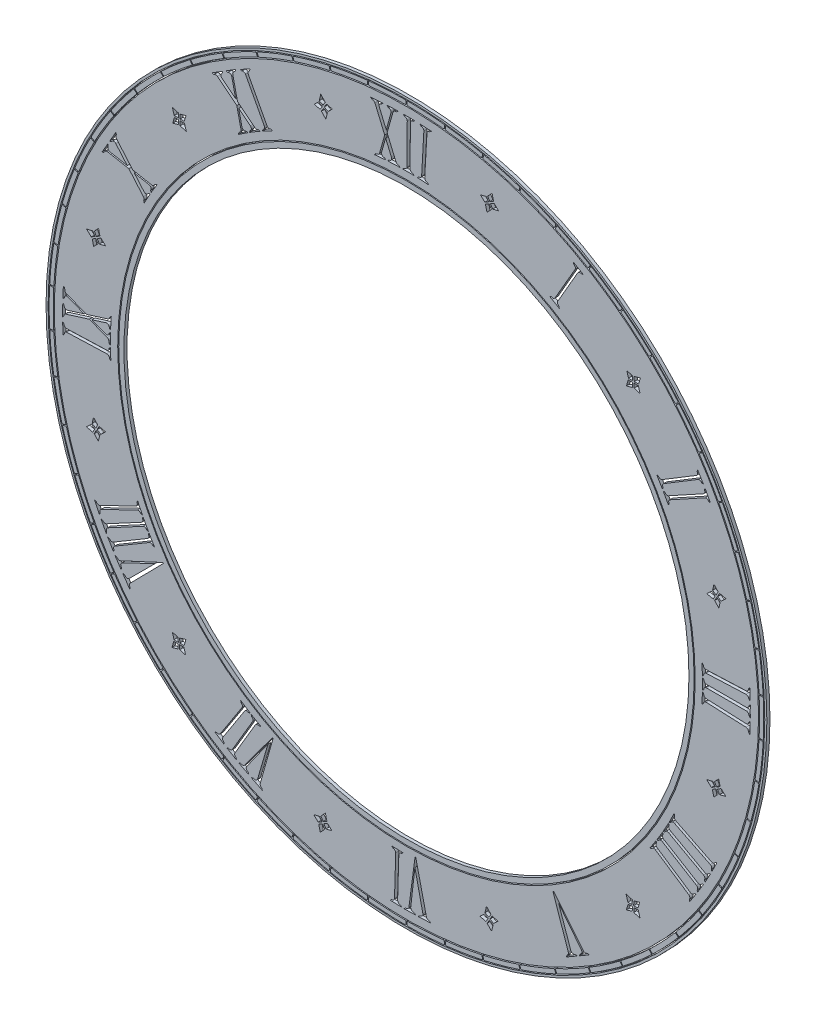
SolidWorks part; units mm, degrees
ref_plane "Спереди" through (0, 0, 0) normal (0, 0, 1) x (1, 0, 0)
ref_plane "Сверху" through (0, 0, 0) normal (0, 1, 0) x (1, 0, 0)
ref_plane "Справа" through (0, 0, 0) normal (1, 0, 0) x (0, 0, -1)
sketch "Эскиз1"
  dimension "D1" = 347
  dimension "D2" = 345
  dimension "D3" = 339
  dimension "D4" = 309.2
  dimension "D8" = 0.745
  dimension "D9" = 0.9
  dimension "D11" = 57
  dimension "D12" = 57
  dimension "D13" = 5
  dimension "D14" = 0.25
  dimension "D15" = 0.083
  dimension "D17" = 170
  dimension "D18" = 5.833
  dimension "D19" = 331
  dimension "D6" = 15
  dimension "D5" = 272
  dimension "D10" = 4.8
  dimension "D16" = 172
  dimension "D20" = 285
  dimension "D22" = 331
  dimension "D23" = 285
  dimension "D26" = 45
  dimension "D27" = 0.635
  dimension "D28" = 2.5
  dimension "D29" = 2.5
  dimension "D31" = 2.5
  dimension "D36" = 2.5
  dimension "D50" = 0.75
  dimension "D52" = 9.5
  dimension "D47" = 5.5
  dimension "D49" = 2.5
  dimension "D46" = 45
  dimension "D48" = 0.635
  dimension "D56" = 2.5
  dimension "D59" = 45
  dimension "D62" = 2.4
  dimension "D74" = 283
  dimension "D75" = 283
  dimension "D76" = 0.365
  dimension "D85" = 9.5
  dimension "D86" = 9.5
  dimension "D88" = 2.5
  dimension "D92" = 45
  dimension "D98" = 1.6
  dimension "D105" = 2.5
  dimension "D118" = 2.5
  dimension "D149" = 11.25
  dimension "D150" = 1.75
  dimension "D145" = 168.998
  dimension "D173" = 6
  dimension "D176" = 9.5
  dimension "D174" = 2.5
  dimension "D192" = 23
  dimension "D163" = 1.25
  dimension "D164" = 1.25
  dimension "D165" = 1.25
  dimension "D166" = 1.25
  dimension "D167" = 5.5
  dimension "D168" = 45
  dimension "D169" = 45
  dimension "D170" = 9.5
  dimension "D179" = 3.5
  dimension "D7" = 1.2
  dimension "D21" = 30
  dimension "D24" = 45
  dimension "D25" = 0.635
  dimension "D30" = 9.5
  dimension "D32" = 9.5
  dimension "D33" = 0.0265
  dimension "D34" = 45
  dimension "D35" = 0.635
  dimension "D37" = 9.5
  dimension "D38" = 2.75
  dimension "D39" = 0.75
  dimension "D40" = 58.8
  dimension "D41" = 30
  dimension "D42" = 30
  dimension "D43" = 30
  dimension "D44" = 0.0265
  dimension "D45" = 0.75
  dimension "D51" = 0.26
  dimension "D53" = 0.0265
  dimension "D54" = 0.75
  dimension "D55" = 2.4
  dimension "D57" = 0.0265
  dimension "D58" = 1.5
  dimension "D60" = 9.5
  dimension "D61" = 0.635
  dimension "D63" = 1.5
  dimension "D64" = 45
  dimension "D65" = 170.5
  dimension "D66" = 45
  dimension "D67" = 170.5
  dimension "D68" = 0.75
  dimension "D69" = 45
  dimension "D70" = 9.5
  dimension "D71" = 5.5
  dimension "D72" = 45
  dimension "D73" = 30
  dimension "D77" = 11.25
  dimension "D78" = 9.25
  dimension "D79" = 0.5
  dimension "D80" = 1
  dimension "D81" = 0.635
  dimension "D82" = 0.365
  dimension "D83" = 45
  dimension "D84" = 45
  dimension "D87" = 5.5
  dimension "D89" = 45
  dimension "D90" = 9.5
  dimension "D91" = 6
  dimension "D93" = 9.5
  dimension "D94" = 2.5
  dimension "D95" = 3.5
  dimension "D96" = 45
  dimension "D97" = 0.635
  dimension "D99" = 1
  dimension "D100" = 0.5
  dimension "D101" = 6
  dimension "D102" = 45
  dimension "D103" = 0.635
  dimension "D104" = 45
  dimension "D106" = 9.5
  dimension "D107" = 9.5
  dimension "D108" = 3.5
  dimension "D109" = 45
  dimension "D110" = 45
  dimension "D111" = 5.5
  dimension "D112" = 3
  dimension "D113" = 9.5
  dimension "D114" = 9.5
  dimension "D115" = 0.5
  dimension "D116" = 11.25
  dimension "D117" = 20.5
  dimension "D119" = 9.5
  dimension "D120" = 0.0265
  dimension "D121" = 1.5
  dimension "D122" = 2.95
  dimension "D123" = 2.4
  dimension "D124" = 2.4
  dimension "D125" = 0.365
  dimension "D126" = 0.5
  dimension "D127" = 1
  dimension "D128" = 0.635
  dimension "D129" = 45
  dimension "D130" = 45
  dimension "D131" = 9.5
  dimension "D132" = 9.5
  dimension "D133" = 5.5
  dimension "D134" = 2.5
  dimension "D135" = 45
  dimension "D136" = 9.5
  dimension "D137" = 6
  dimension "D138" = 45
  dimension "D139" = 9.5
  dimension "D140" = 2.5
  dimension "D141" = 45
  dimension "D142" = 9.5
  dimension "D143" = 0.0265
  dimension "D144" = 1.5
  dimension "D146" = 171.249
  dimension "D147" = 171.249
  dimension "D148" = 168.998
  dimension "D151" = 9.25
  dimension "D152" = 0.5
  dimension "D153" = 1.6
  dimension "D154" = 30
  dimension "D155" = 2.95
  dimension "D156" = 0.365
  dimension "D157" = 0.5
  dimension "D158" = 11.25
  dimension "D159" = 9.25
  dimension "D160" = 0.5
  dimension "D161" = 1
  dimension "D162" = 0.5
  dimension "D171" = 168.998
  dimension "D172" = 45
  dimension "D175" = 30
  dimension "D177" = 9.5
  dimension "D178" = 171.249
  dimension "D194" = 5.251
  dimension "D196" = 14.6674
sketch "Эскиз2" plane through (0, 0, 0) normal (0, 0, 1) x (1, 0, 0)
  line L0 (69.7227, 124.993) -> (70.0277, 124.879) construction
  line L1 (68.8553, 124.7606) -> (69.7227, 124.993) construction
  line L2 (73.3858, 122.8781) -> (73.1345, 123.0853) construction
  line L3 (73.6182, 122.0107) -> (73.3858, 122.8781) construction
  line L4 (72.8471, 124.6748) -> (82.452, 141.311) construction
  line L5 (71.548, 125.4248) -> (81.1529, 142.061) construction
  line L6 (80.6142, 143.8577) -> (80.8655, 143.6506) construction
  line L7 (80.3818, 144.7251) -> (80.6142, 143.8577) construction
  line L8 (84.2773, 141.7428) -> (83.9723, 141.8569) construction
  line L9 (85.1447, 141.9752) -> (84.2773, 141.7428) construction
  line L10 (120.4421, 76.1574) -> (121.3142, 75.9431) construction
  line L11 (121.3142, 75.9431) -> (121.5267, 75.6962) construction
  line L12 (123.2913, 71.4528) -> (123.5055, 72.325) construction
  line L13 (123.5055, 72.325) -> (123.385, 72.6276) construction
  line L14 (140.3303, 84.1102) -> (123.8989, 74.159) construction
  line L15 (139.5533, 85.3933) -> (123.1219, 75.4421) construction
  line L16 (139.9467, 87.2274) -> (140.0672, 86.9247) construction
  line L17 (140.1609, 88.0995) -> (139.9467, 87.2274) construction
  line L18 (142.138, 83.6092) -> (141.9255, 83.8562) construction
  line L19 (143.0101, 83.395) -> (142.138, 83.6092) construction
  line L20 (143.7272, 82.1529) -> (143.4766, 81.2905) construction
  line L21 (143.4766, 81.2905) -> (143.5843, 80.983) construction
  line L22 (143.0068, 79.4745) -> (126.1731, 70.2201) construction
  line L23 (143.7294, 78.16) -> (126.8957, 68.9056) construction
  line L24 (145.5145, 77.5837) -> (145.3126, 77.8394) construction
  line L25 (146.3768, 77.3332) -> (145.5145, 77.5837) construction
  line L26 (123.5256, 71.047) -> (124.388, 70.7964) construction
  line L27 (124.388, 70.7964) -> (124.5899, 70.5408) construction
  line L28 (126.1753, 66.2273) -> (126.4258, 67.0896) construction
  line L29 (126.4258, 67.0896) -> (126.3181, 67.3971) construction
  line L30 (142.8944, 8.1058) -> (142.9615, 7.7871) construction
  line L31 (142.2333, 8.7136) -> (142.8944, 8.1058) construction
  line L32 (143.0715, 3.8797) -> (143.1117, 4.2029) construction
  line L33 (142.4636, 3.2187) -> (143.0715, 3.8797) construction
  line L34 (163.4928, 6.1017) -> (144.2998, 5.2973) construction
  line L35 (163.43, 7.6004) -> (144.237, 6.796) construction
  line L36 (164.6583, 9.018) -> (164.6181, 8.6948) construction
  line L37 (165.2662, 9.679) -> (164.6583, 9.018) construction
  line L38 (164.8355, 4.7919) -> (164.7683, 5.1106) construction
  line L39 (165.4965, 4.1841) -> (164.8355, 4.7919) construction
  line L40 (165.5265, 2.7499) -> (164.8915, 2.1149) construction
  line L41 (164.8915, 2.1149) -> (164.8378, 1.7937) construction
  line L42 (164.8915, -2.1149) -> (164.8378, -1.7937) construction
  line L43 (165.5265, -2.7499) -> (164.8915, -2.1149) construction
  line L44 (163.6049, -0.75) -> (144.3951, -0.75) construction
  line L45 (163.6049, 0.75) -> (144.3951, 0.75) construction
  line L46 (142.4735, 2.7499) -> (143.1085, 2.1149) construction
  line L47 (143.1085, 2.1149) -> (143.1622, 1.7937) construction
  line L48 (142.4735, -2.7499) -> (143.1085, -2.1149) construction
  line L49 (143.1085, -2.1149) -> (143.1622, -1.7937) construction
  line L50 (142.4636, -3.2187) -> (143.0715, -3.8797) construction
  line L51 (143.0715, -3.8797) -> (143.1117, -4.2029) construction
  line L52 (163.4928, -6.1017) -> (144.2998, -5.2973) construction
  line L53 (142.2333, -8.7136) -> (142.8944, -8.1058) construction
  line L54 (142.8944, -8.1058) -> (142.9615, -7.7871) construction
  line L55 (163.43, -7.6004) -> (144.237, -6.796) construction
  line L56 (164.8355, -4.7919) -> (164.7683, -5.1106) construction
  line L57 (165.4965, -4.1841) -> (164.8355, -4.7919) construction
  line L58 (165.2662, -9.679) -> (164.6583, -9.018) construction
  line L59 (164.6583, -9.018) -> (164.6181, -8.6948) construction
  line L60 (126.1753, -66.2273) -> (126.4258, -67.0896) construction
  line L61 (123.5256, -71.047) -> (124.388, -70.7964) construction
  line L62 (124.388, -70.7964) -> (124.5899, -70.5408) construction
  line L63 (143.0068, -79.4745) -> (126.1731, -70.2201) construction
  line L64 (143.7294, -78.16) -> (126.8957, -68.9056) construction
  line L65 (126.4258, -67.0896) -> (126.3181, -67.3971) construction
  line L66 (126.3924, -65.8119) -> (127.2435, -65.5255) construction
  line L67 (127.2435, -65.5255) -> (127.4346, -65.2616) construction
  line L68 (128.8379, -60.8855) -> (129.1243, -61.7366) construction
  line L69 (129.1243, -61.7366) -> (129.0296, -62.0483) construction
  line L70 (146.8763, -72.0727) -> (129.6698, -63.5313) construction
  line L71 (146.2094, -73.4163) -> (129.0029, -64.8749) construction
  line L72 (148.6357, -71.4221) -> (148.4447, -71.686) construction
  line L73 (149.4868, -71.1357) -> (148.6357, -71.4221) construction
  line L74 (146.7549, -75.211) -> (146.8496, -74.8993) construction
  line L75 (147.0413, -76.0621) -> (146.7549, -75.211) construction
  line L76 (145.5145, -77.5837) -> (145.3126, -77.8394) construction
  line L77 (146.3768, -77.3332) -> (145.5145, -77.5837) construction
  line L78 (143.4766, -81.2905) -> (143.5843, -80.983) construction
  line L79 (143.7272, -82.1529) -> (143.4766, -81.2905) construction
  line L80 (123.2913, -71.4528) -> (123.5055, -72.325) construction
  line L81 (123.5055, -72.325) -> (123.385, -72.6276) construction
  line L82 (120.4421, -76.1574) -> (121.3142, -75.9431) construction
  line L83 (121.3142, -75.9431) -> (121.5267, -75.6962) construction
  line L84 (139.5533, -85.3933) -> (123.1219, -75.4421) construction
  line L85 (140.3303, -84.1102) -> (123.8989, -74.159) construction
  line L86 (142.138, -83.6092) -> (141.9255, -83.8562) construction
  line L87 (143.0101, -83.395) -> (142.138, -83.6092) construction
  line L88 (140.1609, -88.0995) -> (139.9467, -87.2274) construction
  line L89 (139.9467, -87.2274) -> (140.0672, -86.9247) construction
  line L90 (138.5121, -89.488) -> (138.2895, -89.7258) construction
  line L91 (139.3924, -89.3105) -> (138.5121, -89.488) construction
  line L92 (136.3487, -93.8915) -> (136.1712, -93.0112) construction
  line L93 (136.1712, -93.0112) -> (136.3043, -92.7138) construction
  line L94 (135.855, -91.1623) -> (119.8547, -80.5317) construction
  line L95 (136.685, -89.9129) -> (120.6848, -79.2823) construction
  line L96 (120.191, -76.5531) -> (120.3685, -77.4334) construction
  line L97 (120.3685, -77.4334) -> (120.2355, -77.7308) construction
  line L98 (118.0276, -80.9566) -> (118.2502, -80.7188) construction
  line L99 (117.1473, -81.1341) -> (118.0276, -80.9566) construction
  line L100 (70.9023, -122.4546) -> (70.5862, -122.6371) construction
  line L101 (70.5862, -122.6371) -> (77.9037, -144.1936) construction
  line L102 (70.9023, -122.4546) -> (85.1495, -139.8923) construction
  line L103 (84.2067, -140.015) -> (73.2913, -126.1689) construction
  line L104 (79.1284, -142.8838) -> (73.2913, -126.1689) construction
  line L105 (77.2397, -145.787) -> (77.5151, -145.56) construction
  line L106 (77.0073, -146.6544) -> (77.2397, -145.787) construction
  line L107 (81.336, -143.422) -> (80.7463, -143.6425) construction
  line L108 (82.2034, -143.6544) -> (81.336, -143.422) construction
  line L109 (83.3171, -143.0088) -> (83.5495, -142.1413) construction
  line L110 (83.5495, -142.1413) -> (84.0202, -141.7534) construction
  line L111 (87.2128, -140.0264) -> (86.5552, -140.2722) construction
  line L112 (88.0802, -140.2588) -> (87.2128, -140.0264) construction
  line L113 (4.1348, -141.4397) -> (4.4996, -141.4286) construction
  line L114 (4.1348, -141.4397) -> (1.1963, -163.7544) construction
  line L115 (4.4996, -141.4286) -> (9.6139, -163.5837) construction
  line L116 (2.0625, -163.3728) -> (4.0666, -145.7872) construction
  line L117 (7.9129, -163.139) -> (4.0666, -145.7872) construction
  line L118 (-0.486, -164.9512) -> (0.1963, -164.8181) construction
  line L119 (-1.1038, -165.6029) -> (-0.486, -164.9512) construction
  line L120 (3.7424, -164.8378) -> (3.1312, -164.7523) construction
  line L121 (4.3942, -165.4556) -> (3.7424, -164.8378) construction
  line L122 (5.6918, -165.4247) -> (6.3025, -164.7662) construction
  line L123 (6.3025, -164.7662) -> (6.945, -164.6337) construction
  line L124 (11.0291, -164.5884) -> (10.672, -164.5423) construction
  line L125 (11.6876, -165.199) -> (11.0291, -164.5884) construction
  line L126 (-7.1496, -164.75) -> (-6.8268, -164.7061) construction
  line L127 (-7.8037, -165.3654) -> (-7.1496, -164.75) construction
  line L128 (-2.3062, -165.5333) -> (-2.9215, -164.8792) construction
  line L129 (-2.9215, -164.8792) -> (-3.241, -164.8157) construction
  line L130 (-4.2466, -163.5515) -> (-3.66, -144.3506) construction
  line L131 (-5.7459, -163.5057) -> (-5.1593, -144.3048) construction
  line L132 (-2.2563, -143.1063) -> (-2.5791, -143.1502) construction
  line L133 (-1.6022, -142.491) -> (-2.2563, -143.1063) construction
  line L134 (-6.4843, -142.9771) -> (-6.1648, -143.0407) construction
  line L135 (-7.0996, -142.323) -> (-6.4843, -142.9771) construction
  line L136 (-79.8876, -144.3159) -> (-80.743, -144.5895) construction
  line L137 (-79.2256, -144.528) -> (-79.8876, -144.3159) construction
  line L138 (-64.5122, -125.9383) -> (-77.8368, -144.0776) construction
  line L139 (-66.6663, -129.7153) -> (-76.894, -144.1605) construction
  line L140 (-76.1275, -146.2536) -> (-76.622, -145.8842) construction
  line L141 (-75.8539, -147.1089) -> (-76.1275, -146.2536) construction
  line L142 (-74.702, -147.7069) -> (-73.8496, -147.4241) construction
  line L143 (-73.8496, -147.4241) -> (-73.2227, -147.6175) construction
  line L144 (-69.6219, -149.5452) -> (-69.9127, -149.3328) construction
  line L145 (-69.3391, -150.3975) -> (-69.6219, -149.5452) construction
  line L146 (-64.1871, -126.1043) -> (-70.3782, -147.983) construction
  line L147 (-66.6663, -129.7153) -> (-71.6545, -146.7739) construction
  line L148 (-64.1871, -126.1043) -> (-64.5122, -125.9383) construction
  line L149 (69.7227, 124.993) -> (70.0277, 124.879)
  line L150 (68.8553, 124.7606) -> (69.7227, 124.993)
  line L151 (73.3858, 122.8781) -> (73.1345, 123.0853)
  line L152 (73.6182, 122.0107) -> (73.3858, 122.8781)
  line L153 (72.8471, 124.6748) -> (82.452, 141.311)
  line L154 (71.548, 125.4248) -> (81.1529, 142.061)
  line L155 (80.6142, 143.8577) -> (80.8655, 143.6506)
  line L156 (80.3818, 144.7251) -> (80.6142, 143.8577)
  line L157 (84.2773, 141.7428) -> (83.9723, 141.8569)
  line L158 (85.1447, 141.9752) -> (84.2773, 141.7428)
  line L159 (120.4421, 76.1574) -> (121.3142, 75.9431)
  line L160 (121.3142, 75.9431) -> (121.5267, 75.6962)
  line L161 (123.2913, 71.4528) -> (123.5055, 72.325)
  line L162 (123.5055, 72.325) -> (123.385, 72.6276)
  line L163 (140.3303, 84.1102) -> (123.8989, 74.159)
  line L164 (139.5533, 85.3933) -> (123.1219, 75.4421)
  line L165 (139.9467, 87.2274) -> (140.0672, 86.9247)
  line L166 (140.1609, 88.0995) -> (139.9467, 87.2274)
  line L167 (142.138, 83.6092) -> (141.9255, 83.8562)
  line L168 (143.0101, 83.395) -> (142.138, 83.6092)
  line L169 (143.7272, 82.1529) -> (143.4766, 81.2905)
  line L170 (143.4766, 81.2905) -> (143.5843, 80.983)
  line L171 (143.0068, 79.4745) -> (126.1731, 70.2201)
  line L172 (143.7294, 78.16) -> (126.8957, 68.9056)
  line L173 (145.5145, 77.5837) -> (145.3126, 77.8394)
  line L174 (146.3768, 77.3332) -> (145.5145, 77.5837)
  line L175 (123.5256, 71.047) -> (124.388, 70.7964)
  line L176 (124.388, 70.7964) -> (124.5899, 70.5408)
  line L177 (126.1753, 66.2273) -> (126.4258, 67.0896)
  line L178 (126.4258, 67.0896) -> (126.3181, 67.3971)
  line L179 (142.8944, 8.1058) -> (142.9615, 7.7871)
  line L180 (142.2333, 8.7136) -> (142.8944, 8.1058)
  line L181 (143.0715, 3.8797) -> (143.1117, 4.2029)
  line L182 (142.4636, 3.2187) -> (143.0715, 3.8797)
  line L183 (163.4928, 6.1017) -> (144.2998, 5.2973)
  line L184 (163.43, 7.6004) -> (144.237, 6.796)
  line L185 (164.6583, 9.018) -> (164.6181, 8.6948)
  line L186 (165.2662, 9.679) -> (164.6583, 9.018)
  line L187 (164.8355, 4.7919) -> (164.7683, 5.1106)
  line L188 (165.4965, 4.1841) -> (164.8355, 4.7919)
  line L189 (165.5265, 2.7499) -> (164.8915, 2.1149)
  line L190 (164.8915, 2.1149) -> (164.8378, 1.7937)
  line L191 (164.8915, -2.1149) -> (164.8378, -1.7937)
  line L192 (165.5265, -2.7499) -> (164.8915, -2.1149)
  line L193 (163.6049, -0.75) -> (144.3951, -0.75)
  line L194 (163.6049, 0.75) -> (144.3951, 0.75)
  line L195 (142.4735, 2.7499) -> (143.1085, 2.1149)
  line L196 (143.1085, 2.1149) -> (143.1622, 1.7937)
  line L197 (142.4735, -2.7499) -> (143.1085, -2.1149)
  line L198 (143.1085, -2.1149) -> (143.1622, -1.7937)
  line L199 (142.4636, -3.2187) -> (143.0715, -3.8797)
  line L200 (143.0715, -3.8797) -> (143.1117, -4.2029)
  line L201 (163.4928, -6.1017) -> (144.2998, -5.2973)
  line L202 (142.2333, -8.7136) -> (142.8944, -8.1058)
  line L203 (142.8944, -8.1058) -> (142.9615, -7.7871)
  line L204 (163.43, -7.6004) -> (144.237, -6.796)
  line L205 (164.8355, -4.7919) -> (164.7683, -5.1106)
  line L206 (165.4965, -4.1841) -> (164.8355, -4.7919)
  line L207 (165.2662, -9.679) -> (164.6583, -9.018)
  line L208 (164.6583, -9.018) -> (164.6181, -8.6948)
  line L209 (126.1753, -66.2273) -> (126.4258, -67.0896)
  line L210 (123.5256, -71.047) -> (124.388, -70.7964)
  line L211 (124.388, -70.7964) -> (124.5899, -70.5408)
  line L212 (143.0068, -79.4745) -> (126.1731, -70.2201)
  line L213 (143.7294, -78.16) -> (126.8957, -68.9056)
  line L214 (126.4258, -67.0896) -> (126.3181, -67.3971)
  line L215 (126.3924, -65.8119) -> (127.2435, -65.5255)
  line L216 (127.2435, -65.5255) -> (127.4346, -65.2616)
  line L217 (128.8379, -60.8855) -> (129.1243, -61.7366)
  line L218 (129.1243, -61.7366) -> (129.0296, -62.0483)
  line L219 (146.8763, -72.0727) -> (129.6698, -63.5313)
  line L220 (146.2094, -73.4163) -> (129.0029, -64.8749)
  line L221 (148.6357, -71.4221) -> (148.4447, -71.686)
  line L222 (149.4868, -71.1357) -> (148.6357, -71.4221)
  line L223 (146.7549, -75.211) -> (146.8496, -74.8993)
  line L224 (147.0413, -76.0621) -> (146.7549, -75.211)
  line L225 (145.5145, -77.5837) -> (145.3126, -77.8394)
  line L226 (146.3768, -77.3332) -> (145.5145, -77.5837)
  line L227 (143.4766, -81.2905) -> (143.5843, -80.983)
  line L228 (143.7272, -82.1529) -> (143.4766, -81.2905)
  line L229 (123.2913, -71.4528) -> (123.5055, -72.325)
  line L230 (123.5055, -72.325) -> (123.385, -72.6276)
  line L231 (120.4421, -76.1574) -> (121.3142, -75.9431)
  line L232 (121.3142, -75.9431) -> (121.5267, -75.6962)
  line L233 (139.5533, -85.3933) -> (123.1219, -75.4421)
  line L234 (140.3303, -84.1102) -> (123.8989, -74.159)
  line L235 (142.138, -83.6092) -> (141.9255, -83.8562)
  line L236 (143.0101, -83.395) -> (142.138, -83.6092)
  line L237 (140.1609, -88.0995) -> (139.9467, -87.2274)
  line L238 (139.9467, -87.2274) -> (140.0672, -86.9247)
  line L239 (138.5121, -89.488) -> (138.2895, -89.7258)
  line L240 (139.3924, -89.3105) -> (138.5121, -89.488)
  line L241 (136.3487, -93.8915) -> (136.1712, -93.0112)
  line L242 (136.1712, -93.0112) -> (136.3043, -92.7138)
  line L243 (135.855, -91.1623) -> (119.8547, -80.5317)
  line L244 (136.685, -89.9129) -> (120.6848, -79.2823)
  line L245 (120.191, -76.5531) -> (120.3685, -77.4334)
  line L246 (120.3685, -77.4334) -> (120.2355, -77.7308)
  line L247 (118.0276, -80.9566) -> (118.2502, -80.7188)
  line L248 (117.1473, -81.1341) -> (118.0276, -80.9566)
  line L249 (70.9023, -122.4546) -> (70.5862, -122.6371)
  line L250 (70.5862, -122.6371) -> (77.9037, -144.1936)
  line L251 (70.9023, -122.4546) -> (85.1495, -139.8923)
  line L252 (84.2067, -140.015) -> (73.2913, -126.1689)
  line L253 (79.1284, -142.8838) -> (73.2913, -126.1689)
  line L254 (77.2397, -145.787) -> (77.5151, -145.56)
  line L255 (77.0073, -146.6544) -> (77.2397, -145.787)
  line L256 (81.336, -143.422) -> (80.7463, -143.6425)
  line L257 (82.2034, -143.6544) -> (81.336, -143.422)
  line L258 (83.3171, -143.0088) -> (83.5495, -142.1413)
  line L259 (83.5495, -142.1413) -> (84.0202, -141.7534)
  line L260 (87.2128, -140.0264) -> (86.5552, -140.2722)
  line L261 (88.0802, -140.2588) -> (87.2128, -140.0264)
  line L262 (4.1348, -141.4397) -> (4.4996, -141.4286)
  line L263 (4.1348, -141.4397) -> (1.1963, -163.7544)
  line L264 (4.4996, -141.4286) -> (9.6139, -163.5837)
  line L265 (2.0625, -163.3728) -> (4.0666, -145.7872)
  line L266 (7.9129, -163.139) -> (4.0666, -145.7872)
  line L267 (-0.486, -164.9512) -> (0.1963, -164.8181)
  line L268 (-1.1038, -165.6029) -> (-0.486, -164.9512)
  line L269 (3.7424, -164.8378) -> (3.1312, -164.7523)
  line L270 (4.3942, -165.4556) -> (3.7424, -164.8378)
  line L271 (5.6918, -165.4247) -> (6.3025, -164.7662)
  line L272 (6.3025, -164.7662) -> (6.945, -164.6337)
  line L273 (11.0291, -164.5884) -> (10.672, -164.5423)
  line L274 (11.6876, -165.199) -> (11.0291, -164.5884)
  line L275 (-7.1496, -164.75) -> (-6.8268, -164.7061)
  line L276 (-7.8037, -165.3654) -> (-7.1496, -164.75)
  line L277 (-2.3062, -165.5333) -> (-2.9215, -164.8792)
  line L278 (-2.9215, -164.8792) -> (-3.241, -164.8157)
  line L279 (-4.2466, -163.5515) -> (-3.66, -144.3506)
  line L280 (-5.7459, -163.5057) -> (-5.1593, -144.3048)
  line L281 (-2.2563, -143.1063) -> (-2.5791, -143.1502)
  line L282 (-1.6022, -142.491) -> (-2.2563, -143.1063)
  line L283 (-6.4843, -142.9771) -> (-6.1648, -143.0407)
  line L284 (-7.0996, -142.323) -> (-6.4843, -142.9771)
  line L285 (-79.8876, -144.3159) -> (-80.743, -144.5895)
  line L286 (-79.2256, -144.528) -> (-79.8876, -144.3159)
  line L287 (-64.5122, -125.9383) -> (-77.8368, -144.0776)
  line L288 (-66.6663, -129.7153) -> (-76.894, -144.1605)
  line L289 (-76.1275, -146.2536) -> (-76.622, -145.8842)
  line L290 (-75.8539, -147.1089) -> (-76.1275, -146.2536)
  line L291 (-74.702, -147.7069) -> (-73.8496, -147.4241)
  line L292 (-73.8496, -147.4241) -> (-73.2227, -147.6175)
  line L293 (-69.6219, -149.5452) -> (-69.9127, -149.3328)
  line L294 (-69.3391, -150.3975) -> (-69.6219, -149.5452)
  line L295 (-64.1871, -126.1043) -> (-70.3782, -147.983)
  line L296 (-66.6663, -129.7153) -> (-71.6545, -146.7739)
  line L297 (-64.1871, -126.1043) -> (-64.5122, -125.9383)
  line L300 (-41.9806, 150.8749) -> (-41.2463, 153.9335) construction
  line L301 (-41.2463, 153.9335) -> (-39.0811, 151.6518) construction
  line L303 (-40.1687, 149.9117) -> (-41.9806, 150.8749) construction
  line L304 (0, 0) -> (0, 173.5) construction
  line L305 (0, 0) -> (0, 173.5) construction
  line L306 (-42.259, 150.1791) -> (-44.3862, 148.1604) construction
  line L307 (0, 0) -> (-41.2463, 153.9335) construction
  line L308 (0, 0) -> (-41.2463, 153.9335) construction
  line L309 (-40.4471, 149.2159) -> (-42.259, 150.1791) construction
  line L310 (-41.5347, 147.4758) -> (-44.3862, 148.1604) construction
  line L311 (-40.4471, 149.2159) -> (-41.5347, 147.4758) construction
  line L312 (-39.8581, 148.7526) -> (-40.9457, 147.0125) construction
  line L313 (-40.9457, 147.0125) -> (-38.7805, 144.7308) construction
  line L314 (-38.7805, 144.7308) -> (-38.0462, 147.7894) construction
  line L315 (-39.8581, 148.7526) -> (-38.0462, 147.7894) construction
  line L316 (-39.5798, 149.4483) -> (-37.7678, 148.4851) construction
  line L317 (-39.5798, 149.4483) -> (-38.4922, 151.1884) construction
  line L318 (-38.4922, 151.1884) -> (-35.6406, 150.5038) construction
  line L319 (-37.7678, 148.4851) -> (-35.6406, 150.5038) construction
  line L320 (-41.9806, 150.8749) -> (-41.2463, 153.9335)
  line L321 (-41.2463, 153.9335) -> (-39.0811, 151.6518)
  line L322 (-40.1687, 149.9117) -> (-41.9806, 150.8749)
  line L323 (-42.259, 150.1791) -> (-44.3862, 148.1604)
  line L324 (-40.4471, 149.2159) -> (-42.259, 150.1791)
  line L325 (-41.5347, 147.4758) -> (-44.3862, 148.1604)
  line L326 (-40.4471, 149.2159) -> (-41.5347, 147.4758)
  line L327 (-39.8581, 148.7526) -> (-40.9457, 147.0125)
  line L328 (-40.9457, 147.0125) -> (-38.7805, 144.7308)
  line L329 (-38.7805, 144.7308) -> (-38.0462, 147.7894)
  line L330 (-39.8581, 148.7526) -> (-38.0462, 147.7894)
  line L331 (-39.5798, 149.4483) -> (-37.7678, 148.4851)
  line L332 (-39.5798, 149.4483) -> (-38.4922, 151.1884)
  line L333 (-38.4922, 151.1884) -> (-35.6406, 150.5038)
  line L334 (-37.7678, 148.4851) -> (-35.6406, 150.5038)
  line L335 (39.064, 151.5878) -> (41.2292, 153.8694)
  line L336 (41.2292, 153.8694) -> (41.9635, 150.8108)
  line L337 (40.1516, 149.8477) -> (39.064, 151.5878)
  line L338 (38.475, 151.1244) -> (35.6234, 150.4398)
  line L339 (39.5626, 149.3843) -> (38.475, 151.1244)
  line L340 (37.7507, 148.4211) -> (35.6234, 150.4398)
  line L341 (39.5626, 149.3843) -> (37.7507, 148.4211)
  line L342 (39.841, 148.6885) -> (38.029, 147.7254)
  line L343 (38.029, 147.7254) -> (38.7633, 144.6668)
  line L344 (38.7633, 144.6668) -> (40.9286, 146.9484)
  line L345 (39.841, 148.6885) -> (40.9286, 146.9484)
  line L346 (40.4299, 149.1519) -> (41.5175, 147.4118)
  line L347 (40.4299, 149.1519) -> (42.2418, 150.1151)
  line L348 (42.2418, 150.1151) -> (44.3691, 148.0964)
  line L349 (41.5175, 147.4118) -> (44.3691, 148.0964)
  line L350 (109.6071, 111.6828) -> (112.6231, 112.5762)
  line L351 (112.6231, 112.5762) -> (111.7297, 109.5602)
  line L352 (109.6789, 109.6321) -> (109.6071, 111.6828)
  line L353 (108.8654, 111.576) -> (106.0535, 112.4089)
  line L354 (108.9372, 109.5252) -> (108.8654, 111.576)
  line L355 (106.8865, 109.5971) -> (106.0535, 112.4089)
  line L356 (108.9372, 109.5252) -> (106.8865, 109.5971)
  line L357 (108.8304, 108.7835) -> (106.7796, 108.8553)
  line L358 (106.7796, 108.8553) -> (105.8863, 105.8394)
  line L359 (105.8863, 105.8394) -> (108.9022, 106.7328)
  line L360 (108.8304, 108.7835) -> (108.9022, 106.7328)
  line L361 (109.5721, 108.8903) -> (109.6439, 106.8396)
  line L362 (109.5721, 108.8903) -> (111.6229, 108.8185)
  line L363 (111.6229, 108.8185) -> (112.4558, 106.0067)
  line L364 (109.6439, 106.8396) -> (112.4558, 106.0067)
  line L365 (150.7468, 41.8526) -> (153.8054, 41.1183)
  line L366 (153.8054, 41.1183) -> (151.5237, 38.9531)
  line L367 (149.7836, 40.0406) -> (150.7468, 41.8526)
  line L368 (150.051, 42.1309) -> (148.0324, 44.2582)
  line L369 (149.0879, 40.319) -> (150.051, 42.1309)
  line L370 (147.3478, 41.4066) -> (148.0324, 44.2582)
  line L371 (149.0879, 40.319) -> (147.3478, 41.4066)
  line L372 (148.6245, 39.7301) -> (146.8844, 40.8176)
  line L373 (146.8844, 40.8176) -> (144.6027, 38.6524)
  line L374 (144.6027, 38.6524) -> (147.6613, 37.9181)
  line L375 (148.6245, 39.7301) -> (147.6613, 37.9181)
  line L376 (149.3203, 39.4517) -> (148.3571, 37.6398)
  line L377 (149.3203, 39.4517) -> (151.0604, 38.3641)
  line L378 (151.0604, 38.3641) -> (150.3758, 35.5125)
  line L379 (148.3571, 37.6398) -> (150.3758, 35.5125)
  line L380 (151.4597, -39.192) -> (153.7413, -41.3573)
  line L381 (153.7413, -41.3573) -> (150.6828, -42.0916)
  line L382 (149.7196, -40.2796) -> (151.4597, -39.192)
  line L383 (150.9963, -38.6031) -> (150.3117, -35.7515)
  line L384 (149.2562, -39.6907) -> (150.9963, -38.6031)
  line L385 (148.293, -37.8788) -> (150.3117, -35.7515)
  line L386 (149.2562, -39.6907) -> (148.293, -37.8788)
  line L387 (148.5605, -39.969) -> (147.5973, -38.1571)
  line L388 (147.5973, -38.1571) -> (144.5387, -38.8914)
  line L389 (144.5387, -38.8914) -> (146.8204, -41.0566)
  line L390 (148.5605, -39.969) -> (146.8204, -41.0566)
  line L391 (149.0238, -40.558) -> (147.2837, -41.6456)
  line L392 (149.0238, -40.558) -> (149.987, -42.3699)
  line L393 (149.987, -42.3699) -> (147.9683, -44.4972)
  line L394 (147.2837, -41.6456) -> (147.9683, -44.4972)
  line L395 (111.5547, -109.7352) -> (112.4481, -112.7511)
  line L396 (112.4481, -112.7511) -> (109.4322, -111.8578)
  line L397 (109.504, -109.807) -> (111.5547, -109.7352)
  line L398 (111.4479, -108.9935) -> (112.2808, -106.1816)
  line L399 (109.3972, -109.0653) -> (111.4479, -108.9935)
  line L400 (109.469, -107.0145) -> (112.2808, -106.1816)
  line L401 (109.3972, -109.0653) -> (109.469, -107.0145)
  line L402 (108.6555, -108.9585) -> (108.7273, -106.9077)
  line L403 (108.7273, -106.9077) -> (105.7113, -106.0143)
  line L404 (105.7113, -106.0143) -> (106.6047, -109.0303)
  line L405 (108.6555, -108.9585) -> (106.6047, -109.0303)
  line L406 (108.7623, -109.7002) -> (106.7115, -109.772)
  line L407 (108.7623, -109.7002) -> (108.6904, -111.751)
  line L408 (108.6904, -111.751) -> (105.8786, -112.5839)
  line L409 (106.7115, -109.772) -> (105.8786, -112.5839)
  line L410 (41.7245, -150.8749) -> (40.9902, -153.9335)
  line L411 (40.9902, -153.9335) -> (38.825, -151.6518)
  line L412 (39.9126, -149.9117) -> (41.7245, -150.8749)
  line L413 (42.0029, -150.1791) -> (44.1301, -148.1604)
  line L414 (40.1909, -149.2159) -> (42.0029, -150.1791)
  line L415 (41.2785, -147.4758) -> (44.1301, -148.1604)
  line L416 (40.1909, -149.2159) -> (41.2785, -147.4758)
  line L417 (39.602, -148.7526) -> (40.6896, -147.0125)
  line L418 (40.6896, -147.0125) -> (38.5244, -144.7308)
  line L419 (38.5244, -144.7308) -> (37.7901, -147.7894)
  line L420 (39.602, -148.7526) -> (37.7901, -147.7894)
  line L421 (39.3236, -149.4483) -> (37.5117, -148.4851)
  line L422 (39.3236, -149.4483) -> (38.236, -151.1884)
  line L423 (38.236, -151.1884) -> (35.3844, -150.5038)
  line L424 (37.5117, -148.4851) -> (35.3844, -150.5038)
  line L425 (-39.3201, -151.5878) -> (-41.4853, -153.8694)
  line L426 (-41.4853, -153.8694) -> (-42.2196, -150.8108)
  line L427 (-40.4077, -149.8477) -> (-39.3201, -151.5878)
  line L428 (-38.7312, -151.1244) -> (-35.8796, -150.4398)
  line L429 (-39.8188, -149.3843) -> (-38.7312, -151.1244)
  line L430 (-38.0068, -148.4211) -> (-35.8796, -150.4398)
  line L431 (-39.8188, -149.3843) -> (-38.0068, -148.4211)
  line L432 (-40.0971, -148.6885) -> (-38.2852, -147.7254)
  line L433 (-38.2852, -147.7254) -> (-39.0195, -144.6668)
  line L434 (-39.0195, -144.6668) -> (-41.1847, -146.9484)
  line L435 (-40.0971, -148.6885) -> (-41.1847, -146.9484)
  line L436 (-40.6861, -149.1519) -> (-41.7736, -147.4118)
  line L437 (-40.6861, -149.1519) -> (-42.498, -150.1151)
  line L438 (-42.498, -150.1151) -> (-44.6252, -148.0964)
  line L439 (-41.7736, -147.4118) -> (-44.6252, -148.0964)
  line L440 (-109.8633, -111.6828) -> (-112.8792, -112.5762)
  line L441 (-112.8792, -112.5762) -> (-111.9859, -109.5602)
  line L442 (-109.9351, -109.6321) -> (-109.8633, -111.6828)
  line L443 (-109.1215, -111.576) -> (-106.3097, -112.4089)
  line L444 (-109.1934, -109.5252) -> (-109.1215, -111.576)
  line L445 (-107.1426, -109.5971) -> (-106.3097, -112.4089)
  line L446 (-109.1934, -109.5252) -> (-107.1426, -109.5971)
  line L447 (-109.0866, -108.7835) -> (-107.0358, -108.8553)
  line L448 (-107.0358, -108.8553) -> (-106.1424, -105.8394)
  line L449 (-106.1424, -105.8394) -> (-109.1584, -106.7328)
  line L450 (-109.0866, -108.7835) -> (-109.1584, -106.7328)
  line L451 (-109.8283, -108.8903) -> (-109.9001, -106.8396)
  line L452 (-109.8283, -108.8903) -> (-111.879, -108.8185)
  line L453 (-111.879, -108.8185) -> (-112.712, -106.0067)
  line L454 (-109.9001, -106.8396) -> (-112.712, -106.0067)
  line L455 (-151.0029, -41.8526) -> (-154.0615, -41.1183)
  line L456 (-154.0615, -41.1183) -> (-151.7799, -38.9531)
  line L457 (-150.0398, -40.0406) -> (-151.0029, -41.8526)
  line L458 (-150.3072, -42.1309) -> (-148.2885, -44.2582)
  line L459 (-149.344, -40.319) -> (-150.3072, -42.1309)
  line L460 (-147.6039, -41.4066) -> (-148.2885, -44.2582)
  line L461 (-149.344, -40.319) -> (-147.6039, -41.4066)
  line L462 (-148.8807, -39.7301) -> (-147.1405, -40.8176)
  line L463 (-147.1405, -40.8176) -> (-144.8589, -38.6524)
  line L464 (-144.8589, -38.6524) -> (-147.9175, -37.9181)
  line L465 (-148.8807, -39.7301) -> (-147.9175, -37.9181)
  line L466 (-149.5764, -39.4517) -> (-148.6132, -37.6398)
  line L467 (-149.5764, -39.4517) -> (-151.3165, -38.3641)
  line L468 (-151.3165, -38.3641) -> (-150.6319, -35.5125)
  line L469 (-148.6132, -37.6398) -> (-150.6319, -35.5125)
  line L470 (-151.7158, 39.192) -> (-153.9975, 41.3573)
  line L471 (-153.9975, 41.3573) -> (-150.9389, 42.0916)
  line L472 (-149.9757, 40.2796) -> (-151.7158, 39.192)
  line L473 (-151.2525, 38.6031) -> (-150.5679, 35.7515)
  line L474 (-149.5124, 39.6907) -> (-151.2525, 38.6031)
  line L475 (-148.5492, 37.8788) -> (-150.5679, 35.7515)
  line L476 (-149.5124, 39.6907) -> (-148.5492, 37.8788)
  line L477 (-148.8166, 39.969) -> (-147.8534, 38.1571)
  line L478 (-147.8534, 38.1571) -> (-144.7949, 38.8914)
  line L479 (-144.7949, 38.8914) -> (-147.0765, 41.0566)
  line L480 (-148.8166, 39.969) -> (-147.0765, 41.0566)
  line L481 (-149.28, 40.558) -> (-147.5399, 41.6456)
  line L482 (-149.28, 40.558) -> (-150.2432, 42.3699)
  line L483 (-150.2432, 42.3699) -> (-148.2245, 44.4972)
  line L484 (-147.5399, 41.6456) -> (-148.2245, 44.4972)
  line L485 (-111.8109, 109.7352) -> (-112.7043, 112.7511)
  line L486 (-112.7043, 112.7511) -> (-109.6883, 111.8578)
  line L487 (-109.7601, 109.807) -> (-111.8109, 109.7352)
  line L488 (-111.7041, 108.9935) -> (-112.537, 106.1816)
  line L489 (-109.6533, 109.0653) -> (-111.7041, 108.9935)
  line L490 (-109.7251, 107.0145) -> (-112.537, 106.1816)
  line L491 (-109.6533, 109.0653) -> (-109.7251, 107.0145)
  line L492 (-108.9116, 108.9585) -> (-108.9834, 106.9077)
  line L493 (-108.9834, 106.9077) -> (-105.9675, 106.0143)
  line L494 (-105.9675, 106.0143) -> (-106.8608, 109.0303)
  line L495 (-108.9116, 108.9585) -> (-106.8608, 109.0303)
  line L496 (-109.0184, 109.7002) -> (-106.9676, 109.772)
  line L497 (-109.0184, 109.7002) -> (-108.9466, 111.751)
  line L498 (-108.9466, 111.751) -> (-106.1347, 112.5839)
  line L499 (-106.9676, 109.772) -> (-106.1347, 112.5839)
  line L500 (-40.1687, 149.9117) -> (-39.0811, 151.6518) construction
  line L501 (-40.1687, 149.9117) -> (-39.0811, 151.6518)
  line L502 (40.1516, 149.8477) -> (41.9635, 150.8108)
  line L503 (109.6789, 109.6321) -> (111.7297, 109.5602)
  line L504 (149.7836, 40.0406) -> (151.5237, 38.9531)
  line L505 (149.7196, -40.2796) -> (150.6828, -42.0916)
  line L506 (109.504, -109.807) -> (109.4322, -111.8578)
  line L507 (39.9126, -149.9117) -> (38.825, -151.6518)
  line L508 (-40.4077, -149.8477) -> (-42.2196, -150.8108)
  line L509 (-109.9351, -109.6321) -> (-111.9859, -109.5602)
  line L510 (-150.0398, -40.0406) -> (-151.7799, -38.9531)
  line L511 (-149.9757, 40.2796) -> (-150.9389, 42.0916)
  line L512 (-109.7601, 109.807) -> (-109.6883, 111.8578)
  circle A0 centre (0, 0) radius 136 construction
  circle A1 centre (0, 0) radius 173.5 construction
  arc A2 (70.0277, 124.879) -> (71.548, 125.4248) centre (70.4655, 126.0498) ccw construction
  arc A3 (73.6182, 122.0107) -> (68.8553, 124.7606) centre (0, 0) ccw construction
  arc A4 (72.8471, 124.6748) -> (73.1345, 123.0853) centre (73.9296, 124.0498) ccw construction
  arc A5 (81.1529, 142.061) -> (80.8655, 143.6506) centre (80.0704, 142.686) ccw construction
  arc A6 (80.3818, 144.7251) -> (85.1447, 141.9752) centre (154, 266.7358) ccw construction
  arc A7 (83.9723, 141.8569) -> (82.452, 141.311) centre (83.5345, 140.686) ccw construction
  arc A8 (123.2913, 71.4528) -> (120.4421, 76.1574) centre (0, 0) ccw construction
  arc A9 (121.5267, 75.6962) -> (123.1219, 75.4421) centre (122.4743, 76.5113) ccw construction
  arc A10 (123.8989, 74.159) -> (123.385, 72.6276) centre (124.5465, 73.0898) ccw construction
  arc A11 (139.5533, 85.3933) -> (140.0672, 86.9247) centre (138.9057, 86.4625) ccw construction
  arc A12 (140.1609, 88.0995) -> (143.0101, 83.395) centre (263.4522, 159.5523) ccw construction
  arc A13 (141.9255, 83.8562) -> (140.3303, 84.1102) centre (140.9778, 83.041) ccw construction
  arc A14 (143.7272, 82.1529) -> (146.3768, 77.3332) centre (269.9025, 148.3801) ccw construction
  arc A15 (143.0068, 79.4745) -> (143.5843, 80.983) centre (142.4046, 80.5699) ccw construction
  arc A16 (145.3126, 77.8394) -> (143.7294, 78.16) centre (144.3316, 77.0647) ccw construction
  arc A17 (126.1753, 66.2273) -> (123.5256, 71.047) centre (0, 0) ccw construction
  arc A18 (124.5899, 70.5408) -> (126.1731, 70.2201) centre (125.5709, 71.3155) ccw construction
  arc A19 (126.8957, 68.9056) -> (126.3181, 67.3971) centre (127.4979, 67.8103) ccw construction
  arc A20 (142.9615, 7.7871) -> (144.237, 6.796) centre (144.1847, 8.0449) ccw construction
  arc A21 (142.4636, 3.2187) -> (142.2333, 8.7136) centre (0, 0) ccw construction
  arc A22 (144.2998, 5.2973) -> (143.1117, 4.2029) centre (144.3522, 4.0484) ccw construction
  arc A23 (163.43, 7.6004) -> (164.6181, 8.6948) centre (163.3777, 8.8493) ccw construction
  arc A24 (164.7683, 5.1106) -> (163.4928, 6.1017) centre (163.5452, 4.8528) ccw construction
  arc A25 (165.2662, 9.679) -> (165.4965, 4.1841) centre (307.7298, 12.8977) ccw construction
  arc A26 (165.5265, 2.7499) -> (165.5265, -2.7499) centre (308, 0) ccw construction
  arc A27 (163.6049, 0.75) -> (164.8378, 1.7937) centre (163.6049, 2) ccw construction
  arc A28 (164.8378, -1.7937) -> (163.6049, -0.75) centre (163.6049, -2) ccw construction
  arc A29 (142.4735, -2.7499) -> (142.4735, 2.7499) centre (0, 0) ccw construction
  arc A30 (143.1622, 1.7937) -> (144.3951, 0.75) centre (144.3951, 2) ccw construction
  arc A31 (144.3951, -0.75) -> (143.1622, -1.7937) centre (144.3951, -2) ccw construction
  arc A32 (142.2333, -8.7136) -> (142.4636, -3.2187) centre (0, 0) ccw construction
  arc A33 (143.1117, -4.2029) -> (144.2998, -5.2973) centre (144.3522, -4.0484) ccw construction
  arc A34 (144.237, -6.796) -> (142.9615, -7.7871) centre (144.1847, -8.0449) ccw construction
  arc A35 (163.4928, -6.1017) -> (164.7683, -5.1106) centre (163.5452, -4.8528) ccw construction
  arc A36 (165.4965, -4.1841) -> (165.2662, -9.679) centre (307.7298, -12.8977) ccw construction
  arc A37 (164.6181, -8.6948) -> (163.43, -7.6004) centre (163.3777, -8.8493) ccw construction
  arc A38 (126.3924, -65.8119) -> (128.8379, -60.8855) centre (0, 0) ccw construction
  arc A39 (123.5256, -71.047) -> (126.1753, -66.2273) centre (0, 0) ccw construction
  arc A40 (126.1731, -70.2201) -> (124.5899, -70.5408) centre (125.5709, -71.3155) ccw construction
  arc A41 (126.3181, -67.3971) -> (126.8957, -68.9056) centre (127.4979, -67.8103) ccw construction
  arc A42 (129.0296, -62.0483) -> (129.6698, -63.5313) centre (130.2256, -62.4117) ccw construction
  arc A43 (129.0029, -64.8749) -> (127.4346, -65.2616) centre (128.4471, -65.9946) ccw construction
  arc A44 (146.8763, -72.0727) -> (148.4447, -71.686) centre (147.4321, -70.9531) ccw construction
  arc A45 (149.4868, -71.1357) -> (147.0413, -76.0621) centre (275.8792, -136.9476) ccw construction
  arc A46 (146.8496, -74.8993) -> (146.2094, -73.4163) centre (145.6536, -74.5359) ccw construction
  arc A47 (143.7294, -78.16) -> (145.3126, -77.8394) centre (144.3316, -77.0647) ccw construction
  arc A48 (143.5843, -80.983) -> (143.0068, -79.4745) centre (142.4046, -80.5699) ccw construction
  arc A49 (146.3768, -77.3332) -> (143.7272, -82.1529) centre (269.9025, -148.3801) ccw construction
  arc A50 (120.4421, -76.1574) -> (123.2913, -71.4528) centre (0, 0) ccw construction
  arc A51 (123.385, -72.6276) -> (123.8989, -74.159) centre (124.5465, -73.0898) ccw construction
  arc A52 (123.1219, -75.4421) -> (121.5267, -75.6962) centre (122.4743, -76.5113) ccw construction
  arc A53 (140.3303, -84.1102) -> (141.9255, -83.8562) centre (140.9778, -83.041) ccw construction
  arc A54 (143.0101, -83.395) -> (140.1609, -88.0995) centre (263.4522, -159.5523) ccw construction
  arc A55 (140.0672, -86.9247) -> (139.5533, -85.3933) centre (138.9057, -86.4625) ccw construction
  arc A56 (136.685, -89.9129) -> (138.2895, -89.7258) centre (137.3768, -88.8717) ccw construction
  arc A57 (139.3924, -89.3105) -> (136.3487, -93.8915) centre (256.5397, -170.4446) ccw construction
  arc A58 (136.3043, -92.7138) -> (135.855, -91.1623) centre (135.1632, -92.2034) ccw construction
  arc A59 (117.1473, -81.1341) -> (120.191, -76.5531) centre (0, 0) ccw construction
  arc A60 (120.2355, -77.7308) -> (120.6848, -79.2823) centre (121.3765, -78.2412) ccw construction
  arc A61 (119.8547, -80.5317) -> (118.2502, -80.7188) centre (119.1629, -81.5729) ccw construction
  arc A62 (77.5151, -145.56) -> (77.9037, -144.1936) centre (76.72, -144.5954) ccw construction
  arc A63 (82.2034, -143.6544) -> (77.0073, -146.6544) centre (150.8396, -268.5357) ccw construction
  arc A64 (79.1284, -142.8838) -> (80.7463, -143.6425) centre (80.3085, -142.4717) ccw construction
  arc A65 (88.0802, -140.2588) -> (83.3171, -143.0088) centre (156.9351, -265.0196) ccw construction
  arc A66 (84.0202, -141.7534) -> (84.2067, -140.015) centre (83.2251, -140.7888) ccw construction
  arc A67 (85.1495, -139.8923) -> (86.5552, -140.2722) centre (86.1175, -139.1014) ccw construction
  arc A68 (-7.0996, -142.323) -> (-1.6022, -142.491) centre (0, 0) ccw construction
  arc A69 (0.1963, -164.8181) -> (1.1963, -163.7544) centre (-0.043, -163.5912) ccw construction
  arc A70 (4.3942, -165.4556) -> (-1.1038, -165.6029) centre (5.4633, -307.9515) ccw construction
  arc A71 (2.0625, -163.3728) -> (3.1312, -164.7523) centre (3.3044, -163.5143) ccw construction
  arc A72 (11.6876, -165.199) -> (5.6918, -165.4247) centre (14.0475, -307.6795) ccw construction
  arc A73 (6.945, -164.6337) -> (7.9129, -163.139) centre (6.6925, -163.4095) ccw construction
  arc A74 (9.6139, -163.5837) -> (10.672, -164.5423) centre (10.8318, -163.3026) ccw construction
  arc A75 (-6.8268, -164.7061) -> (-5.7459, -163.5057) centre (-6.9953, -163.4675) ccw construction
  arc A76 (-2.3062, -165.5333) -> (-7.8037, -165.3654) centre (-9.4059, -307.8563) ccw construction
  arc A77 (-4.2466, -163.5515) -> (-3.241, -164.8157) centre (-2.9972, -163.5897) ccw construction
  arc A78 (-2.5791, -143.1502) -> (-3.66, -144.3506) centre (-2.4105, -144.3888) ccw construction
  arc A79 (-5.1593, -144.3048) -> (-6.1648, -143.0407) centre (-6.4087, -144.2667) ccw construction
  arc A80 (-75.8539, -147.1089) -> (-80.743, -144.5895) centre (-143.5615, -272.4961) ccw construction
  arc A81 (-79.2256, -144.528) -> (-77.8368, -144.0776) centre (-78.8442, -143.3376) ccw construction
  arc A82 (-76.894, -144.1605) -> (-76.622, -145.8842) centre (-75.8738, -144.8828) ccw construction
  arc A83 (-69.3391, -150.3975) -> (-74.702, -147.7069) centre (-135.9079, -276.3929) ccw construction
  arc A84 (-73.2227, -147.6175) -> (-71.6545, -146.7739) centre (-72.8543, -146.423) ccw construction
  arc A85 (-70.3782, -147.983) -> (-69.9127, -149.3328) centre (-69.1754, -148.3234) ccw construction
  circle A86 centre (0, 0) radius 136
  circle A87 centre (0, 0) radius 173.5
  arc A88 (70.0277, 124.879) -> (71.548, 125.4248) centre (70.4655, 126.0498) ccw
  arc A89 (73.6182, 122.0107) -> (68.8553, 124.7606) centre (0, 0) ccw
  arc A90 (72.8471, 124.6748) -> (73.1345, 123.0853) centre (73.9296, 124.0498) ccw
  arc A91 (81.1529, 142.061) -> (80.8655, 143.6506) centre (80.0704, 142.686) ccw
  arc A92 (80.3818, 144.7251) -> (85.1447, 141.9752) centre (154, 266.7358) ccw
  arc A93 (83.9723, 141.8569) -> (82.452, 141.311) centre (83.5345, 140.686) ccw
  arc A94 (123.2913, 71.4528) -> (120.4421, 76.1574) centre (0, 0) ccw
  arc A95 (121.5267, 75.6962) -> (123.1219, 75.4421) centre (122.4743, 76.5113) ccw
  arc A96 (123.8989, 74.159) -> (123.385, 72.6276) centre (124.5465, 73.0898) ccw
  arc A97 (139.5533, 85.3933) -> (140.0672, 86.9247) centre (138.9057, 86.4625) ccw
  arc A98 (140.1609, 88.0995) -> (143.0101, 83.395) centre (263.4522, 159.5523) ccw
  arc A99 (141.9255, 83.8562) -> (140.3303, 84.1102) centre (140.9778, 83.041) ccw
  arc A100 (143.7272, 82.1529) -> (146.3768, 77.3332) centre (269.9025, 148.3801) ccw
  arc A101 (143.0068, 79.4745) -> (143.5843, 80.983) centre (142.4046, 80.5699) ccw
  arc A102 (145.3126, 77.8394) -> (143.7294, 78.16) centre (144.3316, 77.0647) ccw
  arc A103 (126.1753, 66.2273) -> (123.5256, 71.047) centre (0, 0) ccw
  arc A104 (124.5899, 70.5408) -> (126.1731, 70.2201) centre (125.5709, 71.3155) ccw
  arc A105 (126.8957, 68.9056) -> (126.3181, 67.3971) centre (127.4979, 67.8103) ccw
  arc A106 (142.9615, 7.7871) -> (144.237, 6.796) centre (144.1847, 8.0449) ccw
  arc A107 (142.4636, 3.2187) -> (142.2333, 8.7136) centre (0, 0) ccw
  arc A108 (144.2998, 5.2973) -> (143.1117, 4.2029) centre (144.3522, 4.0484) ccw
  arc A109 (163.43, 7.6004) -> (164.6181, 8.6948) centre (163.3777, 8.8493) ccw
  arc A110 (164.7683, 5.1106) -> (163.4928, 6.1017) centre (163.5452, 4.8528) ccw
  arc A111 (165.2662, 9.679) -> (165.4965, 4.1841) centre (307.7298, 12.8977) ccw
  arc A112 (165.5265, 2.7499) -> (165.5265, -2.7499) centre (308, 0) ccw
  arc A113 (163.6049, 0.75) -> (164.8378, 1.7937) centre (163.6049, 2) ccw
  arc A114 (164.8378, -1.7937) -> (163.6049, -0.75) centre (163.6049, -2) ccw
  arc A115 (142.4735, -2.7499) -> (142.4735, 2.7499) centre (0, 0) ccw
  arc A116 (143.1622, 1.7937) -> (144.3951, 0.75) centre (144.3951, 2) ccw
  arc A117 (144.3951, -0.75) -> (143.1622, -1.7937) centre (144.3951, -2) ccw
  arc A118 (142.2333, -8.7136) -> (142.4636, -3.2187) centre (0, 0) ccw
  arc A119 (143.1117, -4.2029) -> (144.2998, -5.2973) centre (144.3522, -4.0484) ccw
  arc A120 (144.237, -6.796) -> (142.9615, -7.7871) centre (144.1847, -8.0449) ccw
  arc A121 (163.4928, -6.1017) -> (164.7683, -5.1106) centre (163.5452, -4.8528) ccw
  arc A122 (165.4965, -4.1841) -> (165.2662, -9.679) centre (307.7298, -12.8977) ccw
  arc A123 (164.6181, -8.6948) -> (163.43, -7.6004) centre (163.3777, -8.8493) ccw
  arc A124 (126.3924, -65.8119) -> (128.8379, -60.8855) centre (0, 0) ccw
  arc A125 (123.5256, -71.047) -> (126.1753, -66.2273) centre (0, 0) ccw
  arc A126 (126.1731, -70.2201) -> (124.5899, -70.5408) centre (125.5709, -71.3155) ccw
  arc A127 (126.3181, -67.3971) -> (126.8957, -68.9056) centre (127.4979, -67.8103) ccw
  arc A128 (129.0296, -62.0483) -> (129.6698, -63.5313) centre (130.2256, -62.4117) ccw
  arc A129 (129.0029, -64.8749) -> (127.4346, -65.2616) centre (128.4471, -65.9946) ccw
  arc A130 (146.8763, -72.0727) -> (148.4447, -71.686) centre (147.4321, -70.9531) ccw
  arc A131 (149.4868, -71.1357) -> (147.0413, -76.0621) centre (275.8792, -136.9476) ccw
  arc A132 (146.8496, -74.8993) -> (146.2094, -73.4163) centre (145.6536, -74.5359) ccw
  arc A133 (143.7294, -78.16) -> (145.3126, -77.8394) centre (144.3316, -77.0647) ccw
  arc A134 (143.5843, -80.983) -> (143.0068, -79.4745) centre (142.4046, -80.5699) ccw
  arc A135 (146.3768, -77.3332) -> (143.7272, -82.1529) centre (269.9025, -148.3801) ccw
  arc A136 (120.4421, -76.1574) -> (123.2913, -71.4528) centre (0, 0) ccw
  arc A137 (123.385, -72.6276) -> (123.8989, -74.159) centre (124.5465, -73.0898) ccw
  arc A138 (123.1219, -75.4421) -> (121.5267, -75.6962) centre (122.4743, -76.5113) ccw
  arc A139 (140.3303, -84.1102) -> (141.9255, -83.8562) centre (140.9778, -83.041) ccw
  arc A140 (143.0101, -83.395) -> (140.1609, -88.0995) centre (263.4522, -159.5523) ccw
  arc A141 (140.0672, -86.9247) -> (139.5533, -85.3933) centre (138.9057, -86.4625) ccw
  arc A142 (136.685, -89.9129) -> (138.2895, -89.7258) centre (137.3768, -88.8717) ccw
  arc A143 (139.3924, -89.3105) -> (136.3487, -93.8915) centre (256.5397, -170.4446) ccw
  arc A144 (136.3043, -92.7138) -> (135.855, -91.1623) centre (135.1632, -92.2034) ccw
  arc A145 (117.1473, -81.1341) -> (120.191, -76.5531) centre (0, 0) ccw
  arc A146 (120.2355, -77.7308) -> (120.6848, -79.2823) centre (121.3765, -78.2412) ccw
  arc A147 (119.8547, -80.5317) -> (118.2502, -80.7188) centre (119.1629, -81.5729) ccw
  arc A148 (77.5151, -145.56) -> (77.9037, -144.1936) centre (76.72, -144.5954) ccw
  arc A149 (82.2034, -143.6544) -> (77.0073, -146.6544) centre (150.8396, -268.5357) ccw
  arc A150 (79.1284, -142.8838) -> (80.7463, -143.6425) centre (80.3085, -142.4717) ccw
  arc A151 (88.0802, -140.2588) -> (83.3171, -143.0088) centre (156.9351, -265.0196) ccw
  arc A152 (84.0202, -141.7534) -> (84.2067, -140.015) centre (83.2251, -140.7888) ccw
  arc A153 (85.1495, -139.8923) -> (86.5552, -140.2722) centre (86.1175, -139.1014) ccw
  arc A154 (-7.0996, -142.323) -> (-1.6022, -142.491) centre (0, 0) ccw
  arc A155 (0.1963, -164.8181) -> (1.1963, -163.7544) centre (-0.043, -163.5912) ccw
  arc A156 (4.3942, -165.4556) -> (-1.1038, -165.6029) centre (5.4633, -307.9515) ccw
  arc A157 (2.0625, -163.3728) -> (3.1312, -164.7523) centre (3.3044, -163.5143) ccw
  arc A158 (11.6876, -165.199) -> (5.6918, -165.4247) centre (14.0475, -307.6795) ccw
  arc A159 (6.945, -164.6337) -> (7.9129, -163.139) centre (6.6925, -163.4095) ccw
  arc A160 (9.6139, -163.5837) -> (10.672, -164.5423) centre (10.8318, -163.3026) ccw
  arc A161 (-6.8268, -164.7061) -> (-5.7459, -163.5057) centre (-6.9953, -163.4675) ccw
  arc A162 (-2.3062, -165.5333) -> (-7.8037, -165.3654) centre (-9.4059, -307.8563) ccw
  arc A163 (-4.2466, -163.5515) -> (-3.241, -164.8157) centre (-2.9972, -163.5897) ccw
  arc A164 (-2.5791, -143.1502) -> (-3.66, -144.3506) centre (-2.4105, -144.3888) ccw
  arc A165 (-5.1593, -144.3048) -> (-6.1648, -143.0407) centre (-6.4087, -144.2667) ccw
  arc A166 (-75.8539, -147.1089) -> (-80.743, -144.5895) centre (-143.5615, -272.4961) ccw
  arc A167 (-79.2256, -144.528) -> (-77.8368, -144.0776) centre (-78.8442, -143.3376) ccw
  arc A168 (-76.894, -144.1605) -> (-76.622, -145.8842) centre (-75.8738, -144.8828) ccw
  arc A169 (-69.3391, -150.3975) -> (-74.702, -147.7069) centre (-135.9079, -276.3929) ccw
  arc A170 (-73.2227, -147.6175) -> (-71.6545, -146.7739) centre (-72.8543, -146.423) ccw
  arc A171 (-70.3782, -147.983) -> (-69.9127, -149.3328) centre (-69.1754, -148.3234) ccw
  circle A178 centre (0, 0) radius 154.6 construction
  circle A184 centre (0, 0) radius 172.5 construction
  circle A185 centre (0, 0) radius 169.5 construction
  circle A186 centre (0, 0) radius 172.5
  circle A187 centre (0, 0) radius 169.5
  dimension "D1" = 12
  dimension "D2" = 12
extrude "Бобышка-Вытянуть1" add sketch "Эскиз2" along normal blind 1.5 contours A187 L280 A165 L283 L284 A154 L282 L281 A164 L279 A163 L278 L277 A162 L276 L275 A161 L251 A153 L260 L261 A151 L258 L259 A152 L252 L253 A150 L256 L257 A149 L255 L254 A148 L250 L249 L238 A141 L233 A138 L232 L231 A136 L229 L230 A137 L234 A139 | A87 A186
sketch "Эскиз4" plane through (0, 0, 0) normal (0, 0, 1) x (1, 0, 0)
  line L3 (0, 173.5) -> (0, -173.5) construction
  line L4 (173.5, 0) -> (-173.5, 0) construction
  line L5 (0, 0) -> (0, 173.5) construction
  line L6 (0, 0) -> (18.7586, 172.4829) construction
  line L7 (0, 0) -> (37.2974, 169.4437) construction
  line L8 (0, 0) -> (55.3988, 164.4178) construction
  line L9 (0, 0) -> (72.8508, 157.4643) construction
  line L10 (0, 0) -> (89.4486, 148.6647) construction
  line L11 (0, 0) -> (104.9977, 138.1221) construction
  line L12 (0, 0) -> (119.3159, 125.9602) construction
  line L13 (0, 0) -> (132.2351, 112.3215) construction
  line L14 (0, 0) -> (143.604, 97.366) construction
  line L15 (0, 0) -> (153.2893, 81.2689) construction
  line L16 (0, 0) -> (161.1775, 64.219) construction
  line L17 (0, 0) -> (167.1759, 46.4162) construction
  line L18 (0, 0) -> (171.2144, 28.0692) construction
  line L19 (0, 0) -> (173.2455, 9.3931) construction
  line L20 (0, 0) -> (173.2455, -9.3931) construction
  line L21 (0, 0) -> (171.2144, -28.0692) construction
  line L22 (0, 0) -> (167.1759, -46.4162) construction
  line L23 (0, 0) -> (161.1775, -64.219) construction
  line L24 (0, 0) -> (153.2893, -81.2689) construction
  line L25 (0, 0) -> (143.604, -97.366) construction
  line L26 (0, 0) -> (132.2351, -112.3215) construction
  line L27 (0, 0) -> (119.3159, -125.9602) construction
  line L28 (0, 0) -> (104.9977, -138.1221) construction
  line L29 (0, 0) -> (89.4486, -148.6647) construction
  line L30 (0, 0) -> (72.8508, -157.4643) construction
  line L31 (0, 0) -> (55.3988, -164.4178) construction
  line L32 (0, 0) -> (37.2974, -169.4437) construction
  line L33 (0, 0) -> (18.7586, -172.4829) construction
  line L34 (0, 0) -> (0, -173.5) construction
  line L35 (0, 0) -> (-18.7586, -172.4829) construction
  line L36 (0, 0) -> (-37.2974, -169.4437) construction
  line L37 (0, 0) -> (-55.3988, -164.4178) construction
  line L38 (0, 0) -> (-72.8508, -157.4643) construction
  line L39 (0, 0) -> (-89.4486, -148.6647) construction
  line L40 (0, 0) -> (-104.9977, -138.1221) construction
  line L41 (0, 0) -> (-119.3159, -125.9602) construction
  line L42 (0, 0) -> (-132.2351, -112.3215) construction
  line L43 (0, 0) -> (-143.604, -97.366) construction
  line L44 (0, 0) -> (-153.2893, -81.2689) construction
  line L45 (0, 0) -> (-161.1775, -64.219) construction
  line L46 (0, 0) -> (-167.1759, -46.4162) construction
  line L47 (0, 0) -> (-171.2144, -28.0692) construction
  line L48 (0, 0) -> (-173.2455, -9.3931) construction
  line L49 (0, 0) -> (-173.2455, 9.3931) construction
  line L50 (0, 0) -> (-171.2144, 28.0692) construction
  line L51 (0, 0) -> (-167.1759, 46.4162) construction
  line L52 (0, 0) -> (-161.1775, 64.219) construction
  line L53 (0, 0) -> (-153.2893, 81.2689) construction
  line L54 (0, 0) -> (-143.604, 97.366) construction
  line L55 (0, 0) -> (-132.2351, 112.3215) construction
  line L56 (0, 0) -> (-119.3159, 125.9602) construction
  line L57 (0, 0) -> (-104.9977, 138.1221) construction
  line L58 (0, 0) -> (-89.4486, 148.6647) construction
  line L59 (0, 0) -> (-72.8508, 157.4643) construction
  line L60 (0, 0) -> (-55.3988, 164.4178) construction
  line L61 (0, 0) -> (-37.2974, 169.4437) construction
  line L62 (0, 0) -> (-18.7586, 172.4829) construction
  line L63 (-0.25, 171.6051) -> (-0.25, 175.6577) construction
  line L64 (-0.25, 170.3988) -> (-0.25, 171.5988)
  line L65 (-18.3046, 170.6199) -> (-18.1748, 169.4269)
  line L66 (18.1748, 169.4269) -> (18.3046, 170.6199)
  line L67 (0.25, 171.5988) -> (0.25, 170.3988)
  line L68 (36.3865, 166.4687) -> (36.6445, 167.6406)
  line L69 (18.8016, 170.5658) -> (18.6719, 169.3728)
  line L70 (54.1717, 161.5588) -> (54.5548, 162.6959)
  line L71 (37.1328, 167.5331) -> (36.8749, 166.3612)
  line L72 (71.3217, 154.7547) -> (71.8256, 155.8438)
  line L73 (55.0287, 162.5363) -> (54.6455, 161.3991)
  line L74 (87.6355, 146.1363) -> (88.2542, 147.1645)
  line L75 (72.2793, 155.6339) -> (71.7755, 154.5448)
  line L76 (102.9219, 135.8046) -> (103.6481, 136.7599)
  line L77 (88.6826, 146.9067) -> (88.064, 145.8785)
  line L78 (117.0016, 123.8807) -> (117.8269, 124.7519)
  line L79 (104.0462, 136.4573) -> (103.32, 135.502)
  line L80 (129.7096, 110.5044) -> (130.6242, 111.2812)
  line L81 (118.1899, 124.408) -> (117.3646, 123.5368)
  line L82 (140.8969, 95.8325) -> (141.8901, 96.5059)
  line L83 (130.9479, 110.9001) -> (130.0333, 110.1233)
  line L84 (150.4323, 80.0371) -> (151.4925, 80.5992)
  line L85 (142.1707, 96.0921) -> (141.1775, 95.4187)
  line L86 (158.2039, 63.3033) -> (159.3187, 63.7475)
  line L87 (151.7267, 80.1574) -> (150.6665, 79.5953)
  line L88 (164.1208, 45.8274) -> (165.2771, 46.1484)
  line L89 (159.5038, 63.283) -> (158.389, 62.8388)
  line L90 (168.1136, 27.8142) -> (169.2978, 28.0083)
  line L91 (165.4109, 45.6666) -> (164.2546, 45.3456)
  line L92 (170.1353, 9.4748) -> (171.3336, 9.5398)
  line L93 (169.3787, 27.5149) -> (168.1945, 27.3207)
  line L94 (170.1624, -8.9756) -> (171.3606, -9.0405)
  line L95 (171.3606, 9.0405) -> (170.1624, 8.9756)
  line L96 (168.1945, -27.3207) -> (169.3787, -27.5149)
  line L97 (171.3336, -9.5398) -> (170.1353, -9.4748)
  line L98 (164.2546, -45.3456) -> (165.4109, -45.6666)
  line L99 (169.2978, -28.0083) -> (168.1136, -27.8142)
  line L100 (158.389, -62.8388) -> (159.5038, -63.283)
  line L101 (165.2771, -46.1484) -> (164.1208, -45.8274)
  line L102 (150.6665, -79.5953) -> (151.7267, -80.1574)
  line L103 (159.3187, -63.7475) -> (158.2039, -63.3033)
  line L104 (141.1775, -95.4187) -> (142.1707, -96.0921)
  line L105 (151.4925, -80.5992) -> (150.4323, -80.0371)
  line L106 (130.0333, -110.1233) -> (130.9479, -110.9001)
  line L107 (141.8901, -96.5059) -> (140.8969, -95.8325)
  line L108 (117.3646, -123.5368) -> (118.1899, -124.408)
  line L109 (130.6242, -111.2812) -> (129.7096, -110.5044)
  line L110 (103.32, -135.502) -> (104.0462, -136.4573)
  line L111 (117.8269, -124.7519) -> (117.0016, -123.8807)
  line L112 (88.064, -145.8785) -> (88.6826, -146.9067)
  line L113 (103.6481, -136.7599) -> (102.9219, -135.8046)
  line L114 (71.7755, -154.5448) -> (72.2793, -155.6339)
  line L115 (88.2542, -147.1645) -> (87.6355, -146.1363)
  line L116 (54.6455, -161.3991) -> (55.0287, -162.5363)
  line L117 (71.8256, -155.8438) -> (71.3217, -154.7547)
  line L118 (36.8749, -166.3612) -> (37.1328, -167.5331)
  line L119 (54.5548, -162.6959) -> (54.1717, -161.5588)
  line L120 (18.6719, -169.3728) -> (18.8016, -170.5658)
  line L121 (36.6445, -167.6406) -> (36.3865, -166.4687)
  line L122 (0.25, -170.3988) -> (0.25, -171.5988)
  line L123 (18.3046, -170.6199) -> (18.1748, -169.4269)
  line L124 (-18.1748, -169.4269) -> (-18.3046, -170.6199)
  line L125 (-0.25, -171.5988) -> (-0.25, -170.3988)
  line L126 (-36.3865, -166.4687) -> (-36.6445, -167.6406)
  line L127 (-18.8016, -170.5658) -> (-18.6719, -169.3728)
  line L128 (-54.1717, -161.5588) -> (-54.5548, -162.6959)
  line L129 (-37.1328, -167.5331) -> (-36.8749, -166.3612)
  line L130 (-71.3217, -154.7547) -> (-71.8256, -155.8438)
  line L131 (-55.0287, -162.5363) -> (-54.6455, -161.3991)
  line L132 (-87.6355, -146.1363) -> (-88.2542, -147.1645)
  line L133 (-72.2793, -155.6339) -> (-71.7755, -154.5448)
  line L134 (-102.9219, -135.8046) -> (-103.6481, -136.7599)
  line L135 (-88.6826, -146.9067) -> (-88.064, -145.8785)
  line L136 (-117.0016, -123.8807) -> (-117.8269, -124.7519)
  line L137 (-104.0462, -136.4573) -> (-103.32, -135.502)
  line L138 (-129.7096, -110.5044) -> (-130.6242, -111.2812)
  line L139 (-118.1899, -124.408) -> (-117.3646, -123.5368)
  line L140 (-140.8969, -95.8325) -> (-141.8901, -96.5059)
  line L141 (-130.9479, -110.9001) -> (-130.0333, -110.1233)
  line L142 (-150.4323, -80.0371) -> (-151.4925, -80.5992)
  line L143 (-142.1707, -96.0921) -> (-141.1775, -95.4187)
  line L144 (-158.2039, -63.3033) -> (-159.3187, -63.7475)
  line L145 (-151.7267, -80.1574) -> (-150.6665, -79.5953)
  line L146 (-164.1208, -45.8274) -> (-165.2771, -46.1484)
  line L147 (-159.5038, -63.283) -> (-158.389, -62.8388)
  line L148 (-168.1136, -27.8142) -> (-169.2978, -28.0083)
  line L149 (-165.4109, -45.6666) -> (-164.2546, -45.3456)
  line L150 (-170.1353, -9.4748) -> (-171.3336, -9.5398)
  line L151 (-169.3787, -27.5149) -> (-168.1945, -27.3207)
  line L152 (-170.1624, 8.9756) -> (-171.3606, 9.0405)
  line L153 (-171.3606, -9.0405) -> (-170.1624, -8.9756)
  line L154 (-168.1945, 27.3207) -> (-169.3787, 27.5149)
  line L155 (-171.3336, 9.5398) -> (-170.1353, 9.4748)
  line L156 (-164.2546, 45.3456) -> (-165.4109, 45.6666)
  line L157 (-169.2978, 28.0083) -> (-168.1136, 27.8142)
  line L158 (-158.389, 62.8388) -> (-159.5038, 63.283)
  line L159 (-165.2771, 46.1484) -> (-164.1208, 45.8274)
  line L160 (-150.6665, 79.5953) -> (-151.7267, 80.1574)
  line L161 (-159.3187, 63.7475) -> (-158.2039, 63.3033)
  line L162 (-141.1775, 95.4187) -> (-142.1707, 96.0921)
  line L163 (-151.4925, 80.5992) -> (-150.4323, 80.0371)
  line L164 (-130.0333, 110.1233) -> (-130.9479, 110.9001)
  line L165 (-141.8901, 96.5059) -> (-140.8969, 95.8325)
  line L166 (-117.3646, 123.5368) -> (-118.1899, 124.408)
  line L167 (-130.6242, 111.2812) -> (-129.7096, 110.5044)
  line L168 (-103.32, 135.502) -> (-104.0462, 136.4573)
  line L169 (-117.8269, 124.7519) -> (-117.0016, 123.8807)
  line L170 (-88.064, 145.8785) -> (-88.6826, 146.9067)
  line L171 (-103.6481, 136.7599) -> (-102.9219, 135.8046)
  line L172 (-71.7755, 154.5448) -> (-72.2793, 155.6339)
  line L173 (-88.2542, 147.1645) -> (-87.6355, 146.1363)
  line L174 (-54.6455, 161.3991) -> (-55.0287, 162.5363)
  line L175 (-71.8256, 155.8438) -> (-71.3217, 154.7547)
  line L176 (-36.8749, 166.3612) -> (-37.1328, 167.5331)
  line L177 (-54.5548, 162.6959) -> (-54.1717, 161.5588)
  line L178 (-18.6719, 169.3728) -> (-18.8016, 170.5658)
  line L179 (-36.6445, 167.6406) -> (-36.3865, 166.4687)
  circle A0 centre (0, 0) radius 173.5 construction
  circle A1 centre (0, 0) radius 173.5 construction
  arc A4 (-0.641, 169.9988) -> (-17.5246, 169.0943) centre (0, 0) ccw construction
  arc A5 (-0.6458, 171.9988) -> (-17.7308, 171.0837) centre (0, 0) ccw construction
  arc A6 (-0.6485, 169.9988) -> (-17.7354, 169.0723) centre (0, 0) ccw
  arc A7 (-0.6515, 171.9988) -> (-17.9486, 171.0609) centre (0, 0) ccw
  arc A8 (-17.7354, 169.0723) -> (-18.1748, 169.4269) centre (-17.7772, 169.4702) cw
  arc A9 (-17.9486, 171.0609) -> (-18.3046, 170.6199) centre (-17.9069, 170.6631) ccw
  arc A10 (-0.6485, 169.9988) -> (-0.25, 170.3988) centre (-0.65, 170.3988) ccw
  arc A11 (-0.6515, 171.9988) -> (-0.25, 171.5988) centre (-0.65, 171.5988) cw
  arc A12 (17.7354, 169.0723) -> (0.6485, 169.9988) centre (0, 0) ccw
  arc A13 (17.9486, 171.0609) -> (0.6515, 171.9988) centre (0, 0) ccw
  arc A14 (0.6485, 169.9988) -> (0.25, 170.3988) centre (0.65, 170.3988) cw
  arc A15 (0.6515, 171.9988) -> (0.25, 171.5988) centre (0.65, 171.5988) ccw
  arc A16 (17.7354, 169.0723) -> (18.1748, 169.4269) centre (17.7772, 169.4702) ccw
  arc A17 (17.9486, 171.0609) -> (18.3046, 170.6199) centre (17.9069, 170.6631) cw
  arc A18 (35.9114, 166.1637) -> (19.0248, 168.9321) centre (0, 0) ccw
  arc A19 (36.3384, 168.1176) -> (19.244, 170.9201) centre (0, 0) ccw
  arc A20 (19.0248, 168.9321) -> (18.6719, 169.3728) centre (19.0695, 169.3296) cw
  arc A21 (19.244, 170.9201) -> (18.8016, 170.5658) centre (19.1993, 170.5226) ccw
  arc A22 (35.9114, 166.1637) -> (36.3865, 166.4687) centre (35.9959, 166.5547) ccw
  arc A23 (36.3384, 168.1176) -> (36.6445, 167.6406) centre (36.2539, 167.7266) cw
  arc A24 (53.6663, 161.3069) -> (37.178, 165.8849) centre (0, 0) ccw
  arc A25 (54.3021, 163.2032) -> (37.6109, 167.8375) centre (0, 0) ccw
  arc A26 (37.178, 165.8849) -> (36.8749, 166.3612) centre (37.2655, 166.2752) cw
  arc A27 (37.6109, 167.8375) -> (37.1328, 167.5331) centre (37.5235, 167.4472) ccw
  arc A28 (53.6663, 161.3069) -> (54.1717, 161.5588) centre (53.7926, 161.6865) ccw
  arc A29 (54.3021, 163.2032) -> (54.5548, 162.6959) centre (54.1758, 162.8237) cw
  arc A30 (70.7921, 154.559) -> (54.8954, 160.8928) centre (0, 0) ccw
  arc A31 (71.6291, 156.3754) -> (55.5369, 162.7871) centre (0, 0) ccw
  arc A32 (54.8954, 160.8928) -> (54.6455, 161.3991) centre (55.0246, 161.2714) cw
  arc A33 (55.5369, 162.7871) -> (55.0287, 162.5363) centre (55.4077, 162.4086) ccw
  arc A34 (70.7921, 154.559) -> (71.3217, 154.7547) centre (70.9587, 154.9227) ccw
  arc A35 (71.6291, 156.3754) -> (71.8256, 155.8438) centre (71.4625, 156.0118) cw
  arc A36 (87.0879, 145.999) -> (71.9692, 154.0144) centre (0, 0) ccw
  arc A37 (88.1164, 147.7143) -> (72.8117, 155.8283) centre (0, 0) ccw
  arc A38 (71.9692, 154.0144) -> (71.7755, 154.5448) centre (72.1385, 154.3768) cw
  arc A39 (72.8117, 155.8283) -> (72.2793, 155.6339) centre (72.6424, 155.4659) ccw
  arc A40 (87.0879, 145.999) -> (87.6355, 146.1363) centre (87.2928, 146.3425) ccw
  arc A41 (88.1164, 147.7143) -> (88.2542, 147.1645) centre (87.9115, 147.3707) cw
  arc A42 (102.3626, 135.7273) -> (88.1992, 145.3303) centre (0, 0) ccw
  arc A43 (103.5706, 137.3213) -> (89.2329, 147.0425) centre (0, 0) ccw
  arc A44 (88.1992, 145.3303) -> (88.064, 145.8785) centre (88.4067, 145.6723) cw
  arc A45 (89.2329, 147.0425) -> (88.6826, 146.9067) centre (89.0254, 146.7005) ccw
  arc A46 (102.3626, 135.7273) -> (102.9219, 135.8046) centre (102.6035, 136.0466) ccw
  arc A47 (103.5706, 137.3213) -> (103.6481, 136.7599) centre (103.3297, 137.002) cw
  arc A48 (116.4373, 123.8643) -> (103.3951, 134.9424) centre (0, 0) ccw
  arc A49 (117.8105, 125.3184) -> (104.6079, 136.5327) centre (0, 0) ccw
  arc A50 (103.3951, 134.9424) -> (103.32, 135.502) centre (103.6384, 135.2599) cw
  arc A51 (104.6079, 136.5327) -> (104.0462, 136.4573) centre (104.3646, 136.2152) ccw
  arc A52 (116.4373, 123.8643) -> (117.0016, 123.8807) centre (116.7112, 124.1557) ccw
  arc A53 (117.8105, 125.3184) -> (117.8269, 124.7519) centre (117.5365, 125.0269) cw
  arc A54 (129.1468, 110.5491) -> (117.3788, 122.9724) centre (0, 0) ccw
  arc A55 (130.6692, 111.8462) -> (118.7565, 124.4223) centre (0, 0) ccw
  arc A56 (117.3788, 122.9724) -> (117.3646, 123.5368) centre (117.655, 123.2617) cw
  arc A57 (118.7565, 124.4223) -> (118.1899, 124.408) centre (118.4803, 124.1329) ccw
  arc A58 (129.1468, 110.5491) -> (129.7096, 110.5044) centre (129.4507, 110.8092) ccw
  arc A59 (130.6692, 111.8462) -> (130.6242, 111.2812) centre (130.3653, 111.5861) cw
  arc A60 (140.3422, 95.9378) -> (129.9864, 109.5606) centre (0, 0) ccw
  arc A61 (141.9959, 97.0627) -> (131.5127, 110.8531) centre (0, 0) ccw
  arc A62 (129.9864, 109.5606) -> (130.0333, 110.1233) centre (130.2923, 109.8184) cw
  arc A63 (131.5127, 110.8531) -> (130.9479, 110.9001) centre (131.2069, 110.5953) ccw
  arc A64 (140.3422, 95.9378) -> (140.8969, 95.8325) centre (140.6724, 96.1636) ccw
  arc A65 (141.9959, 97.0627) -> (141.8901, 96.5059) centre (141.6656, 96.837) cw
  arc A66 (149.8922, 80.2018) -> (141.07, 94.8644) centre (0, 0) ccw
  arc A67 (151.6578, 81.1413) -> (142.7271, 95.9842) centre (0, 0) ccw
  arc A68 (141.07, 94.8644) -> (141.1775, 95.4187) centre (141.402, 95.0876) cw
  arc A69 (142.7271, 95.9842) -> (142.1707, 96.0921) centre (142.3952, 95.761) ccw
  arc A70 (149.8922, 80.2018) -> (150.4323, 80.0371) centre (150.2449, 80.3905) ccw
  arc A71 (151.6578, 81.1413) -> (151.4925, 80.5992) centre (151.3051, 80.9526) cw
  arc A72 (157.6849, 63.5254) -> (150.4997, 79.0559) centre (0, 0) ccw
  arc A73 (159.5417, 64.2685) -> (152.2682, 79.9901) centre (0, 0) ccw
  arc A74 (150.4997, 79.0559) -> (150.6665, 79.5953) centre (150.8538, 79.2419) cw
  arc A75 (152.2682, 79.9901) -> (151.7267, 80.1574) centre (151.914, 79.804) ccw
  arc A76 (157.6849, 63.5254) -> (158.2039, 63.3033) centre (158.0559, 63.6749) ccw
  arc A77 (159.5417, 64.2685) -> (159.3187, 63.7475) centre (159.1707, 64.1191) cw
  arc A78 (163.6288, 46.1043) -> (158.1649, 62.3206) centre (0, 0) ccw
  arc A79 (165.5551, 46.6423) -> (160.024, 63.0581) centre (0, 0) ccw
  arc A80 (158.1649, 62.3206) -> (158.389, 62.8388) centre (158.5371, 62.4672) cw
  arc A81 (160.024, 63.0581) -> (159.5038, 63.283) centre (159.6519, 62.9114) ccw
  arc A82 (163.6288, 46.1043) -> (164.1208, 45.8274) centre (164.0138, 46.2128) ccw
  arc A83 (165.5551, 46.6423) -> (165.2771, 46.1484) centre (165.1701, 46.5338) cw
  arc A84 (167.6544, 28.1427) -> (163.9758, 44.8546) centre (0, 0) ccw
  arc A85 (169.6275, 28.4692) -> (165.9037, 45.3868) centre (0, 0) ccw
  arc A86 (163.9758, 44.8546) -> (164.2546, 45.3456) centre (164.3616, 44.9602) cw
  arc A87 (165.9037, 45.3868) -> (165.4109, 45.6666) centre (165.5179, 45.2812) ccw
  arc A88 (167.6544, 28.1427) -> (168.1136, 27.8142) centre (168.0489, 28.2089) ccw
  arc A89 (169.6275, 28.4692) -> (169.2978, 28.0083) centre (169.2331, 28.403) cw
  arc A90 (169.7143, 9.8511) -> (167.8642, 26.8628) centre (0, 0) ccw
  arc A91 (171.7112, 9.9624) -> (169.8383, 27.1834) centre (0, 0) ccw
  arc A92 (167.8642, 26.8628) -> (168.1945, 27.3207) centre (168.2592, 26.926) cw
  arc A93 (169.8383, 27.1834) -> (169.3787, 27.5149) centre (169.4434, 27.1202) ccw
  arc A94 (169.7143, 9.8511) -> (170.1353, 9.4748) centre (170.1137, 9.8742) ccw
  arc A95 (171.7112, 9.9624) -> (171.3336, 9.5398) centre (171.3119, 9.9392) cw
  arc A96 (169.7846, -8.556) -> (169.7846, 8.556) centre (0, 0) ccw
  arc A97 (171.7818, -8.6613) -> (171.7818, 8.6613) centre (0, 0) ccw
  arc A98 (169.7846, 8.556) -> (170.1624, 8.9756) centre (170.184, 8.5762) cw
  arc A99 (171.7818, 8.6613) -> (171.3606, 9.0405) centre (171.3823, 8.6411) ccw
  arc A100 (169.7846, -8.556) -> (170.1624, -8.9756) centre (170.184, -8.5762) ccw
  arc A101 (171.7818, -8.6613) -> (171.3606, -9.0405) centre (171.3823, -8.6411) cw
  arc A102 (167.8642, -26.8628) -> (169.7143, -9.8511) centre (0, 0) ccw
  arc A103 (169.8383, -27.1834) -> (171.7112, -9.9624) centre (0, 0) ccw
  arc A104 (169.7143, -9.8511) -> (170.1353, -9.4748) centre (170.1137, -9.8742) cw
  arc A105 (171.7112, -9.9624) -> (171.3336, -9.5398) centre (171.3119, -9.9392) ccw
  arc A106 (167.8642, -26.8628) -> (168.1945, -27.3207) centre (168.2592, -26.926) ccw
  arc A107 (169.8383, -27.1834) -> (169.3787, -27.5149) centre (169.4434, -27.1202) cw
  arc A108 (163.9758, -44.8546) -> (167.6544, -28.1427) centre (0, 0) ccw
  arc A109 (165.9037, -45.3868) -> (169.6275, -28.4692) centre (0, 0) ccw
  arc A110 (167.6544, -28.1427) -> (168.1136, -27.8142) centre (168.0489, -28.2089) cw
  arc A111 (169.6275, -28.4692) -> (169.2978, -28.0083) centre (169.2331, -28.403) ccw
  arc A112 (163.9758, -44.8546) -> (164.2546, -45.3456) centre (164.3616, -44.9602) ccw
  arc A113 (165.9037, -45.3868) -> (165.4109, -45.6666) centre (165.5179, -45.2812) cw
  arc A114 (158.1649, -62.3206) -> (163.6288, -46.1043) centre (0, 0) ccw
  arc A115 (160.024, -63.0581) -> (165.5551, -46.6423) centre (0, 0) ccw
  arc A116 (163.6288, -46.1043) -> (164.1208, -45.8274) centre (164.0138, -46.2128) cw
  arc A117 (165.5551, -46.6423) -> (165.2771, -46.1484) centre (165.1701, -46.5338) ccw
  arc A118 (158.1649, -62.3206) -> (158.389, -62.8388) centre (158.5371, -62.4672) ccw
  arc A119 (160.024, -63.0581) -> (159.5038, -63.283) centre (159.6519, -62.9114) cw
  arc A120 (150.4997, -79.0559) -> (157.6849, -63.5254) centre (0, 0) ccw
  arc A121 (152.2682, -79.9901) -> (159.5417, -64.2685) centre (0, 0) ccw
  arc A122 (157.6849, -63.5254) -> (158.2039, -63.3033) centre (158.0559, -63.6749) cw
  arc A123 (159.5417, -64.2685) -> (159.3187, -63.7475) centre (159.1707, -64.1191) ccw
  arc A124 (150.4997, -79.0559) -> (150.6665, -79.5953) centre (150.8538, -79.2419) ccw
  arc A125 (152.2682, -79.9901) -> (151.7267, -80.1574) centre (151.914, -79.804) cw
  arc A126 (141.07, -94.8644) -> (149.8922, -80.2018) centre (0, 0) ccw
  arc A127 (142.7271, -95.9842) -> (151.6578, -81.1413) centre (0, 0) ccw
  arc A128 (149.8922, -80.2018) -> (150.4323, -80.0371) centre (150.2449, -80.3905) cw
  arc A129 (151.6578, -81.1413) -> (151.4925, -80.5992) centre (151.3051, -80.9526) ccw
  arc A130 (141.07, -94.8644) -> (141.1775, -95.4187) centre (141.402, -95.0876) ccw
  arc A131 (142.7271, -95.9842) -> (142.1707, -96.0921) centre (142.3952, -95.761) cw
  arc A132 (129.9864, -109.5606) -> (140.3422, -95.9378) centre (0, 0) ccw
  arc A133 (131.5127, -110.8531) -> (141.9959, -97.0627) centre (0, 0) ccw
  arc A134 (140.3422, -95.9378) -> (140.8969, -95.8325) centre (140.6724, -96.1636) cw
  arc A135 (141.9959, -97.0627) -> (141.8901, -96.5059) centre (141.6656, -96.837) ccw
  arc A136 (129.9864, -109.5606) -> (130.0333, -110.1233) centre (130.2923, -109.8184) ccw
  arc A137 (131.5127, -110.8531) -> (130.9479, -110.9001) centre (131.2069, -110.5953) cw
  arc A138 (117.3788, -122.9724) -> (129.1468, -110.5491) centre (0, 0) ccw
  arc A139 (118.7565, -124.4223) -> (130.6692, -111.8462) centre (0, 0) ccw
  arc A140 (129.1468, -110.5491) -> (129.7096, -110.5044) centre (129.4507, -110.8092) cw
  arc A141 (130.6692, -111.8462) -> (130.6242, -111.2812) centre (130.3653, -111.5861) ccw
  arc A142 (117.3788, -122.9724) -> (117.3646, -123.5368) centre (117.655, -123.2617) ccw
  arc A143 (118.7565, -124.4223) -> (118.1899, -124.408) centre (118.4803, -124.1329) cw
  arc A144 (103.3951, -134.9424) -> (116.4373, -123.8643) centre (0, 0) ccw
  arc A145 (104.6079, -136.5327) -> (117.8105, -125.3184) centre (0, 0) ccw
  arc A146 (116.4373, -123.8643) -> (117.0016, -123.8807) centre (116.7112, -124.1557) cw
  arc A147 (117.8105, -125.3184) -> (117.8269, -124.7519) centre (117.5365, -125.0269) ccw
  arc A148 (103.3951, -134.9424) -> (103.32, -135.502) centre (103.6384, -135.2599) ccw
  arc A149 (104.6079, -136.5327) -> (104.0462, -136.4573) centre (104.3646, -136.2152) cw
  arc A150 (88.1992, -145.3303) -> (102.3626, -135.7273) centre (0, 0) ccw
  arc A151 (89.2329, -147.0425) -> (103.5706, -137.3213) centre (0, 0) ccw
  arc A152 (102.3626, -135.7273) -> (102.9219, -135.8046) centre (102.6035, -136.0466) cw
  arc A153 (103.5706, -137.3213) -> (103.6481, -136.7599) centre (103.3297, -137.002) ccw
  arc A154 (88.1992, -145.3303) -> (88.064, -145.8785) centre (88.4067, -145.6723) ccw
  arc A155 (89.2329, -147.0425) -> (88.6826, -146.9067) centre (89.0254, -146.7005) cw
  arc A156 (71.9692, -154.0144) -> (87.0879, -145.999) centre (0, 0) ccw
  arc A157 (72.8117, -155.8283) -> (88.1164, -147.7143) centre (0, 0) ccw
  arc A158 (87.0879, -145.999) -> (87.6355, -146.1363) centre (87.2928, -146.3425) cw
  arc A159 (88.1164, -147.7143) -> (88.2542, -147.1645) centre (87.9115, -147.3707) ccw
  arc A160 (71.9692, -154.0144) -> (71.7755, -154.5448) centre (72.1385, -154.3768) ccw
  arc A161 (72.8117, -155.8283) -> (72.2793, -155.6339) centre (72.6424, -155.4659) cw
  arc A162 (54.8954, -160.8928) -> (70.7921, -154.559) centre (0, 0) ccw
  arc A163 (55.5369, -162.7871) -> (71.6291, -156.3754) centre (0, 0) ccw
  arc A164 (70.7921, -154.559) -> (71.3217, -154.7547) centre (70.9587, -154.9227) cw
  arc A165 (71.6291, -156.3754) -> (71.8256, -155.8438) centre (71.4625, -156.0118) ccw
  arc A166 (54.8954, -160.8928) -> (54.6455, -161.3991) centre (55.0246, -161.2714) ccw
  arc A167 (55.5369, -162.7871) -> (55.0287, -162.5363) centre (55.4077, -162.4086) cw
  arc A168 (37.178, -165.8849) -> (53.6663, -161.3069) centre (0, 0) ccw
  arc A169 (37.6109, -167.8375) -> (54.3021, -163.2032) centre (0, 0) ccw
  arc A170 (53.6663, -161.3069) -> (54.1717, -161.5588) centre (53.7926, -161.6865) cw
  arc A171 (54.3021, -163.2032) -> (54.5548, -162.6959) centre (54.1758, -162.8237) ccw
  arc A172 (37.178, -165.8849) -> (36.8749, -166.3612) centre (37.2655, -166.2752) ccw
  arc A173 (37.6109, -167.8375) -> (37.1328, -167.5331) centre (37.5235, -167.4472) cw
  arc A174 (19.0248, -168.9321) -> (35.9114, -166.1637) centre (0, 0) ccw
  arc A175 (19.244, -170.9201) -> (36.3384, -168.1176) centre (0, 0) ccw
  arc A176 (35.9114, -166.1637) -> (36.3865, -166.4687) centre (35.9959, -166.5547) cw
  arc A177 (36.3384, -168.1176) -> (36.6445, -167.6406) centre (36.2539, -167.7266) ccw
  arc A178 (19.0248, -168.9321) -> (18.6719, -169.3728) centre (19.0695, -169.3296) ccw
  arc A179 (19.244, -170.9201) -> (18.8016, -170.5658) centre (19.1993, -170.5226) cw
  arc A180 (0.6485, -169.9988) -> (17.7354, -169.0723) centre (0, 0) ccw
  arc A181 (0.6515, -171.9988) -> (17.9486, -171.0609) centre (0, 0) ccw
  arc A182 (17.7354, -169.0723) -> (18.1748, -169.4269) centre (17.7772, -169.4702) cw
  arc A183 (17.9486, -171.0609) -> (18.3046, -170.6199) centre (17.9069, -170.6631) ccw
  arc A184 (0.6485, -169.9988) -> (0.25, -170.3988) centre (0.65, -170.3988) ccw
  arc A185 (0.6515, -171.9988) -> (0.25, -171.5988) centre (0.65, -171.5988) cw
  arc A186 (-17.7354, -169.0723) -> (-0.6485, -169.9988) centre (0, 0) ccw
  arc A187 (-17.9486, -171.0609) -> (-0.6515, -171.9988) centre (0, 0) ccw
  arc A188 (-0.6485, -169.9988) -> (-0.25, -170.3988) centre (-0.65, -170.3988) cw
  arc A189 (-0.6515, -171.9988) -> (-0.25, -171.5988) centre (-0.65, -171.5988) ccw
  arc A190 (-17.7354, -169.0723) -> (-18.1748, -169.4269) centre (-17.7772, -169.4702) ccw
  arc A191 (-17.9486, -171.0609) -> (-18.3046, -170.6199) centre (-17.9069, -170.6631) cw
  arc A192 (-35.9114, -166.1637) -> (-19.0248, -168.9321) centre (0, 0) ccw
  arc A193 (-36.3384, -168.1176) -> (-19.244, -170.9201) centre (0, 0) ccw
  arc A194 (-19.0248, -168.9321) -> (-18.6719, -169.3728) centre (-19.0695, -169.3296) cw
  arc A195 (-19.244, -170.9201) -> (-18.8016, -170.5658) centre (-19.1993, -170.5226) ccw
  arc A196 (-35.9114, -166.1637) -> (-36.3865, -166.4687) centre (-35.9959, -166.5547) ccw
  arc A197 (-36.3384, -168.1176) -> (-36.6445, -167.6406) centre (-36.2539, -167.7266) cw
  arc A198 (-53.6663, -161.3069) -> (-37.178, -165.8849) centre (0, 0) ccw
  arc A199 (-54.3021, -163.2032) -> (-37.6109, -167.8375) centre (0, 0) ccw
  arc A200 (-37.178, -165.8849) -> (-36.8749, -166.3612) centre (-37.2655, -166.2752) cw
  arc A201 (-37.6109, -167.8375) -> (-37.1328, -167.5331) centre (-37.5235, -167.4472) ccw
  arc A202 (-53.6663, -161.3069) -> (-54.1717, -161.5588) centre (-53.7926, -161.6865) ccw
  arc A203 (-54.3021, -163.2032) -> (-54.5548, -162.6959) centre (-54.1758, -162.8237) cw
  arc A204 (-70.7921, -154.559) -> (-54.8954, -160.8928) centre (0, 0) ccw
  arc A205 (-71.6291, -156.3754) -> (-55.5369, -162.7871) centre (0, 0) ccw
  arc A206 (-54.8954, -160.8928) -> (-54.6455, -161.3991) centre (-55.0246, -161.2714) cw
  arc A207 (-55.5369, -162.7871) -> (-55.0287, -162.5363) centre (-55.4077, -162.4086) ccw
  arc A208 (-70.7921, -154.559) -> (-71.3217, -154.7547) centre (-70.9587, -154.9227) ccw
  arc A209 (-71.6291, -156.3754) -> (-71.8256, -155.8438) centre (-71.4625, -156.0118) cw
  arc A210 (-87.0879, -145.999) -> (-71.9692, -154.0144) centre (0, 0) ccw
  arc A211 (-88.1164, -147.7143) -> (-72.8117, -155.8283) centre (0, 0) ccw
  arc A212 (-71.9692, -154.0144) -> (-71.7755, -154.5448) centre (-72.1385, -154.3768) cw
  arc A213 (-72.8117, -155.8283) -> (-72.2793, -155.6339) centre (-72.6424, -155.4659) ccw
  arc A214 (-87.0879, -145.999) -> (-87.6355, -146.1363) centre (-87.2928, -146.3425) ccw
  arc A215 (-88.1164, -147.7143) -> (-88.2542, -147.1645) centre (-87.9115, -147.3707) cw
  arc A216 (-102.3626, -135.7273) -> (-88.1992, -145.3303) centre (0, 0) ccw
  arc A217 (-103.5706, -137.3213) -> (-89.2329, -147.0425) centre (0, 0) ccw
  arc A218 (-88.1992, -145.3303) -> (-88.064, -145.8785) centre (-88.4067, -145.6723) cw
  arc A219 (-89.2329, -147.0425) -> (-88.6826, -146.9067) centre (-89.0254, -146.7005) ccw
  arc A220 (-102.3626, -135.7273) -> (-102.9219, -135.8046) centre (-102.6035, -136.0466) ccw
  arc A221 (-103.5706, -137.3213) -> (-103.6481, -136.7599) centre (-103.3297, -137.002) cw
  arc A222 (-116.4373, -123.8643) -> (-103.3951, -134.9424) centre (0, 0) ccw
  arc A223 (-117.8105, -125.3184) -> (-104.6079, -136.5327) centre (0, 0) ccw
  arc A224 (-103.3951, -134.9424) -> (-103.32, -135.502) centre (-103.6384, -135.2599) cw
  arc A225 (-104.6079, -136.5327) -> (-104.0462, -136.4573) centre (-104.3646, -136.2152) ccw
  arc A226 (-116.4373, -123.8643) -> (-117.0016, -123.8807) centre (-116.7112, -124.1557) ccw
  arc A227 (-117.8105, -125.3184) -> (-117.8269, -124.7519) centre (-117.5365, -125.0269) cw
  arc A228 (-129.1468, -110.5491) -> (-117.3788, -122.9724) centre (0, 0) ccw
  arc A229 (-130.6692, -111.8462) -> (-118.7565, -124.4223) centre (0, 0) ccw
  arc A230 (-117.3788, -122.9724) -> (-117.3646, -123.5368) centre (-117.655, -123.2617) cw
  arc A231 (-118.7565, -124.4223) -> (-118.1899, -124.408) centre (-118.4803, -124.1329) ccw
  arc A232 (-129.1468, -110.5491) -> (-129.7096, -110.5044) centre (-129.4507, -110.8092) ccw
  arc A233 (-130.6692, -111.8462) -> (-130.6242, -111.2812) centre (-130.3653, -111.5861) cw
  arc A234 (-140.3422, -95.9378) -> (-129.9864, -109.5606) centre (0, 0) ccw
  arc A235 (-141.9959, -97.0627) -> (-131.5127, -110.8531) centre (0, 0) ccw
  arc A236 (-129.9864, -109.5606) -> (-130.0333, -110.1233) centre (-130.2923, -109.8184) cw
  arc A237 (-131.5127, -110.8531) -> (-130.9479, -110.9001) centre (-131.2069, -110.5953) ccw
  arc A238 (-140.3422, -95.9378) -> (-140.8969, -95.8325) centre (-140.6724, -96.1636) ccw
  arc A239 (-141.9959, -97.0627) -> (-141.8901, -96.5059) centre (-141.6656, -96.837) cw
  arc A240 (-149.8922, -80.2018) -> (-141.07, -94.8644) centre (0, 0) ccw
  arc A241 (-151.6578, -81.1413) -> (-142.7271, -95.9842) centre (0, 0) ccw
  arc A242 (-141.07, -94.8644) -> (-141.1775, -95.4187) centre (-141.402, -95.0876) cw
  arc A243 (-142.7271, -95.9842) -> (-142.1707, -96.0921) centre (-142.3952, -95.761) ccw
  arc A244 (-149.8922, -80.2018) -> (-150.4323, -80.0371) centre (-150.2449, -80.3905) ccw
  arc A245 (-151.6578, -81.1413) -> (-151.4925, -80.5992) centre (-151.3051, -80.9526) cw
  arc A246 (-157.6849, -63.5254) -> (-150.4997, -79.0559) centre (0, 0) ccw
  arc A247 (-159.5417, -64.2685) -> (-152.2682, -79.9901) centre (0, 0) ccw
  arc A248 (-150.4997, -79.0559) -> (-150.6665, -79.5953) centre (-150.8538, -79.2419) cw
  arc A249 (-152.2682, -79.9901) -> (-151.7267, -80.1574) centre (-151.914, -79.804) ccw
  arc A250 (-157.6849, -63.5254) -> (-158.2039, -63.3033) centre (-158.0559, -63.6749) ccw
  arc A251 (-159.5417, -64.2685) -> (-159.3187, -63.7475) centre (-159.1707, -64.1191) cw
  arc A252 (-163.6288, -46.1043) -> (-158.1649, -62.3206) centre (0, 0) ccw
  arc A253 (-165.5551, -46.6423) -> (-160.024, -63.0581) centre (0, 0) ccw
  arc A254 (-158.1649, -62.3206) -> (-158.389, -62.8388) centre (-158.5371, -62.4672) cw
  arc A255 (-160.024, -63.0581) -> (-159.5038, -63.283) centre (-159.6519, -62.9114) ccw
  arc A256 (-163.6288, -46.1043) -> (-164.1208, -45.8274) centre (-164.0138, -46.2128) ccw
  arc A257 (-165.5551, -46.6423) -> (-165.2771, -46.1484) centre (-165.1701, -46.5338) cw
  arc A258 (-167.6544, -28.1427) -> (-163.9758, -44.8546) centre (0, 0) ccw
  arc A259 (-169.6275, -28.4692) -> (-165.9037, -45.3868) centre (0, 0) ccw
  arc A260 (-163.9758, -44.8546) -> (-164.2546, -45.3456) centre (-164.3616, -44.9602) cw
  arc A261 (-165.9037, -45.3868) -> (-165.4109, -45.6666) centre (-165.5179, -45.2812) ccw
  arc A262 (-167.6544, -28.1427) -> (-168.1136, -27.8142) centre (-168.0489, -28.2089) ccw
  arc A263 (-169.6275, -28.4692) -> (-169.2978, -28.0083) centre (-169.2331, -28.403) cw
  arc A264 (-169.7143, -9.8511) -> (-167.8642, -26.8628) centre (0, 0) ccw
  arc A265 (-171.7112, -9.9624) -> (-169.8383, -27.1834) centre (0, 0) ccw
  arc A266 (-167.8642, -26.8628) -> (-168.1945, -27.3207) centre (-168.2592, -26.926) cw
  arc A267 (-169.8383, -27.1834) -> (-169.3787, -27.5149) centre (-169.4434, -27.1202) ccw
  arc A268 (-169.7143, -9.8511) -> (-170.1353, -9.4748) centre (-170.1137, -9.8742) ccw
  arc A269 (-171.7112, -9.9624) -> (-171.3336, -9.5398) centre (-171.3119, -9.9392) cw
  arc A270 (-169.7846, 8.556) -> (-169.7846, -8.556) centre (0, 0) ccw
  arc A271 (-171.7818, 8.6613) -> (-171.7818, -8.6613) centre (0, 0) ccw
  arc A272 (-169.7846, -8.556) -> (-170.1624, -8.9756) centre (-170.184, -8.5762) cw
  arc A273 (-171.7818, -8.6613) -> (-171.3606, -9.0405) centre (-171.3823, -8.6411) ccw
  arc A274 (-169.7846, 8.556) -> (-170.1624, 8.9756) centre (-170.184, 8.5762) ccw
  arc A275 (-171.7818, 8.6613) -> (-171.3606, 9.0405) centre (-171.3823, 8.6411) cw
  arc A276 (-167.8642, 26.8628) -> (-169.7143, 9.8511) centre (0, 0) ccw
  arc A277 (-169.8383, 27.1834) -> (-171.7112, 9.9624) centre (0, 0) ccw
  arc A278 (-169.7143, 9.8511) -> (-170.1353, 9.4748) centre (-170.1137, 9.8742) cw
  arc A279 (-171.7112, 9.9624) -> (-171.3336, 9.5398) centre (-171.3119, 9.9392) ccw
  arc A280 (-167.8642, 26.8628) -> (-168.1945, 27.3207) centre (-168.2592, 26.926) ccw
  arc A281 (-169.8383, 27.1834) -> (-169.3787, 27.5149) centre (-169.4434, 27.1202) cw
  arc A282 (-163.9758, 44.8546) -> (-167.6544, 28.1427) centre (0, 0) ccw
  arc A283 (-165.9037, 45.3868) -> (-169.6275, 28.4692) centre (0, 0) ccw
  arc A284 (-167.6544, 28.1427) -> (-168.1136, 27.8142) centre (-168.0489, 28.2089) cw
  arc A285 (-169.6275, 28.4692) -> (-169.2978, 28.0083) centre (-169.2331, 28.403) ccw
  arc A286 (-163.9758, 44.8546) -> (-164.2546, 45.3456) centre (-164.3616, 44.9602) ccw
  arc A287 (-165.9037, 45.3868) -> (-165.4109, 45.6666) centre (-165.5179, 45.2812) cw
  arc A288 (-158.1649, 62.3206) -> (-163.6288, 46.1043) centre (0, 0) ccw
  arc A289 (-160.024, 63.0581) -> (-165.5551, 46.6423) centre (0, 0) ccw
  arc A290 (-163.6288, 46.1043) -> (-164.1208, 45.8274) centre (-164.0138, 46.2128) cw
  arc A291 (-165.5551, 46.6423) -> (-165.2771, 46.1484) centre (-165.1701, 46.5338) ccw
  arc A292 (-158.1649, 62.3206) -> (-158.389, 62.8388) centre (-158.5371, 62.4672) ccw
  arc A293 (-160.024, 63.0581) -> (-159.5038, 63.283) centre (-159.6519, 62.9114) cw
  arc A294 (-150.4997, 79.0559) -> (-157.6849, 63.5254) centre (0, 0) ccw
  arc A295 (-152.2682, 79.9901) -> (-159.5417, 64.2685) centre (0, 0) ccw
  arc A296 (-157.6849, 63.5254) -> (-158.2039, 63.3033) centre (-158.0559, 63.6749) cw
  arc A297 (-159.5417, 64.2685) -> (-159.3187, 63.7475) centre (-159.1707, 64.1191) ccw
  arc A298 (-150.4997, 79.0559) -> (-150.6665, 79.5953) centre (-150.8538, 79.2419) ccw
  arc A299 (-152.2682, 79.9901) -> (-151.7267, 80.1574) centre (-151.914, 79.804) cw
  arc A300 (-141.07, 94.8644) -> (-149.8922, 80.2018) centre (0, 0) ccw
  arc A301 (-142.7271, 95.9842) -> (-151.6578, 81.1413) centre (0, 0) ccw
  arc A302 (-149.8922, 80.2018) -> (-150.4323, 80.0371) centre (-150.2449, 80.3905) cw
  arc A303 (-151.6578, 81.1413) -> (-151.4925, 80.5992) centre (-151.3051, 80.9526) ccw
  arc A304 (-141.07, 94.8644) -> (-141.1775, 95.4187) centre (-141.402, 95.0876) ccw
  arc A305 (-142.7271, 95.9842) -> (-142.1707, 96.0921) centre (-142.3952, 95.761) cw
  arc A306 (-129.9864, 109.5606) -> (-140.3422, 95.9378) centre (0, 0) ccw
  arc A307 (-131.5127, 110.8531) -> (-141.9959, 97.0627) centre (0, 0) ccw
  arc A308 (-140.3422, 95.9378) -> (-140.8969, 95.8325) centre (-140.6724, 96.1636) cw
  arc A309 (-141.9959, 97.0627) -> (-141.8901, 96.5059) centre (-141.6656, 96.837) ccw
  arc A310 (-129.9864, 109.5606) -> (-130.0333, 110.1233) centre (-130.2923, 109.8184) ccw
  arc A311 (-131.5127, 110.8531) -> (-130.9479, 110.9001) centre (-131.2069, 110.5953) cw
  arc A312 (-117.3788, 122.9724) -> (-129.1468, 110.5491) centre (0, 0) ccw
  arc A313 (-118.7565, 124.4223) -> (-130.6692, 111.8462) centre (0, 0) ccw
  arc A314 (-129.1468, 110.5491) -> (-129.7096, 110.5044) centre (-129.4507, 110.8092) cw
  arc A315 (-130.6692, 111.8462) -> (-130.6242, 111.2812) centre (-130.3653, 111.5861) ccw
  arc A316 (-117.3788, 122.9724) -> (-117.3646, 123.5368) centre (-117.655, 123.2617) ccw
  arc A317 (-118.7565, 124.4223) -> (-118.1899, 124.408) centre (-118.4803, 124.1329) cw
  arc A318 (-103.3951, 134.9424) -> (-116.4373, 123.8643) centre (0, 0) ccw
  arc A319 (-104.6079, 136.5327) -> (-117.8105, 125.3184) centre (0, 0) ccw
  arc A320 (-116.4373, 123.8643) -> (-117.0016, 123.8807) centre (-116.7112, 124.1557) cw
  arc A321 (-117.8105, 125.3184) -> (-117.8269, 124.7519) centre (-117.5365, 125.0269) ccw
  arc A322 (-103.3951, 134.9424) -> (-103.32, 135.502) centre (-103.6384, 135.2599) ccw
  arc A323 (-104.6079, 136.5327) -> (-104.0462, 136.4573) centre (-104.3646, 136.2152) cw
  arc A324 (-88.1992, 145.3303) -> (-102.3626, 135.7273) centre (0, 0) ccw
  arc A325 (-89.2329, 147.0425) -> (-103.5706, 137.3213) centre (0, 0) ccw
  arc A326 (-102.3626, 135.7273) -> (-102.9219, 135.8046) centre (-102.6035, 136.0466) cw
  arc A327 (-103.5706, 137.3213) -> (-103.6481, 136.7599) centre (-103.3297, 137.002) ccw
  arc A328 (-88.1992, 145.3303) -> (-88.064, 145.8785) centre (-88.4067, 145.6723) ccw
  arc A329 (-89.2329, 147.0425) -> (-88.6826, 146.9067) centre (-89.0254, 146.7005) cw
  arc A330 (-71.9692, 154.0144) -> (-87.0879, 145.999) centre (0, 0) ccw
  arc A331 (-72.8117, 155.8283) -> (-88.1164, 147.7143) centre (0, 0) ccw
  arc A332 (-87.0879, 145.999) -> (-87.6355, 146.1363) centre (-87.2928, 146.3425) cw
  arc A333 (-88.1164, 147.7143) -> (-88.2542, 147.1645) centre (-87.9115, 147.3707) ccw
  arc A334 (-71.9692, 154.0144) -> (-71.7755, 154.5448) centre (-72.1385, 154.3768) ccw
  arc A335 (-72.8117, 155.8283) -> (-72.2793, 155.6339) centre (-72.6424, 155.4659) cw
  arc A336 (-54.8954, 160.8928) -> (-70.7921, 154.559) centre (0, 0) ccw
  arc A337 (-55.5369, 162.7871) -> (-71.6291, 156.3754) centre (0, 0) ccw
  arc A338 (-70.7921, 154.559) -> (-71.3217, 154.7547) centre (-70.9587, 154.9227) cw
  arc A339 (-71.6291, 156.3754) -> (-71.8256, 155.8438) centre (-71.4625, 156.0118) ccw
  arc A340 (-54.8954, 160.8928) -> (-54.6455, 161.3991) centre (-55.0246, 161.2714) ccw
  arc A341 (-55.5369, 162.7871) -> (-55.0287, 162.5363) centre (-55.4077, 162.4086) cw
  arc A342 (-37.178, 165.8849) -> (-53.6663, 161.3069) centre (0, 0) ccw
  arc A343 (-37.6109, 167.8375) -> (-54.3021, 163.2032) centre (0, 0) ccw
  arc A344 (-53.6663, 161.3069) -> (-54.1717, 161.5588) centre (-53.7926, 161.6865) cw
  arc A345 (-54.3021, 163.2032) -> (-54.5548, 162.6959) centre (-54.1758, 162.8237) ccw
  arc A346 (-37.178, 165.8849) -> (-36.8749, 166.3612) centre (-37.2655, 166.2752) ccw
  arc A347 (-37.6109, 167.8375) -> (-37.1328, 167.5331) centre (-37.5235, 167.4472) cw
  arc A348 (-19.0248, 168.9321) -> (-35.9114, 166.1637) centre (0, 0) ccw
  arc A349 (-19.244, 170.9201) -> (-36.3384, 168.1176) centre (0, 0) ccw
  arc A350 (-35.9114, 166.1637) -> (-36.3865, 166.4687) centre (-35.9959, 166.5547) cw
  arc A351 (-36.3384, 168.1176) -> (-36.6445, 167.6406) centre (-36.2539, 167.7266) ccw
  arc A352 (-19.0248, 168.9321) -> (-18.6719, 169.3728) centre (-19.0695, 169.3296) ccw
  arc A353 (-19.244, 170.9201) -> (-18.8016, 170.5658) centre (-19.1993, 170.5226) cw
  dimension "D4" = 0.4
  dimension "D1" = 58
  dimension "D2" = 0.25
  dimension "D3" = 0.25
  dimension "D5" = 58
extrude "Бобышка-Вытянуть2" add sketch "Эскиз4" along normal blind 1.5 separate body
sketch "Эскиз5" plane through (0, 0, 0) normal (0, 0, 1) x (1, 0, 0)
  line L0 (0, -490.6215) -> (0, -325.1215) construction
  line L1 (0, -490.6215) -> (0, -325.1215) construction
  line L2 (0, -490.6215) -> (10.1035, -325.4302) construction
  line L3 (0, -490.6215) -> (10.1035, -325.4302) construction
  line L4 (0, -490.6215) -> (17.0122, -325.9982) construction
  line L5 (0, -490.6215) -> (17.0122, -325.9982) construction
  line L7 (0, 0) -> (-84.122, -142.5263) construction
  line L9 (0, 0) -> (-75.2641, -147.396) construction
  line L10 (-4.3517, -142.4335) -> (-5.0541, -165.4228) construction
  line L11 (-4.3517, -142.4335) -> (-5.0541, -165.4228) construction
  line L12 (-7.0996, -142.323) -> (-6.4843, -142.9771) construction
  line L13 (-6.4843, -142.9771) -> (-6.1648, -143.0407) construction
  line L14 (-1.6022, -142.491) -> (-2.2563, -143.1063) construction
  line L15 (-2.2563, -143.1063) -> (-2.5791, -143.1502) construction
  line L16 (-4.2466, -163.5515) -> (-3.66, -144.3506) construction
  line L17 (-5.7459, -163.5057) -> (-5.1593, -144.3048) construction
  line L18 (-7.1496, -164.75) -> (-6.8268, -164.7061) construction
  line L19 (-7.8037, -165.3654) -> (-7.1496, -164.75) construction
  line L20 (-2.9215, -164.8792) -> (-3.241, -164.8157) construction
  line L21 (-2.3062, -165.5333) -> (-2.9215, -164.8792) construction
  line L22 (-7.0996, -142.323) -> (-6.4843, -142.9771) construction
  line L23 (-6.4843, -142.9771) -> (-6.1648, -143.0407) construction
  line L24 (-1.6022, -142.491) -> (-2.2563, -143.1063) construction
  line L25 (-2.2563, -143.1063) -> (-2.5791, -143.1502) construction
  line L26 (-4.2466, -163.5515) -> (-3.66, -144.3506) construction
  line L27 (-5.7459, -163.5057) -> (-5.1593, -144.3048) construction
  line L28 (-7.1496, -164.75) -> (-6.8268, -164.7061) construction
  line L29 (-7.8037, -165.3654) -> (-7.1496, -164.75) construction
  line L30 (-2.9215, -164.8792) -> (-3.241, -164.8157) construction
  line L31 (-2.3062, -165.5333) -> (-2.9215, -164.8792) construction
  line L32 (-74.7861, -121.2983) -> (-74.562, -122.168)
  line L33 (-74.562, -122.168) -> (-74.3126, -122.3776)
  line L34 (-70.0496, -124.0939) -> (-70.9192, -124.318)
  line L35 (-70.9192, -124.318) -> (-71.2232, -124.201)
  line L36 (-82.5129, -141.2755) -> (-72.7487, -124.7322)
  line L37 (-83.8046, -140.513) -> (-74.0405, -123.9698)
  line L38 (-85.6341, -140.9272) -> (-85.3301, -141.0443)
  line L39 (-86.5038, -141.1513) -> (-85.6341, -140.9272)
  line L40 (-81.9913, -143.0773) -> (-82.2407, -142.8677)
  line L41 (-81.7672, -143.9469) -> (-81.9913, -143.0773)
  line L42 (-72.4313, -122.719) -> (-84.122, -142.5263) construction
  line L43 (-79.8, -118.0602) -> (-79.6125, -118.9385)
  line L44 (-79.6125, -118.9385) -> (-79.3721, -119.1583)
  line L45 (-75.1847, -121.0517) -> (-76.0629, -121.2392)
  line L46 (-76.0629, -121.2392) -> (-76.3618, -121.1095)
  line L47 (-88.3565, -137.6963) -> (-77.9081, -121.5764)
  line L48 (-89.6152, -136.8804) -> (-79.1669, -120.7606)
  line L49 (-91.4604, -137.2176) -> (-91.1616, -137.3473)
  line L50 (-92.3387, -137.4051) -> (-91.4604, -137.2176)
  line L51 (-87.9109, -139.5184) -> (-88.1512, -139.2985)
  line L52 (-87.7234, -140.3966) -> (-87.9109, -139.5184)
  line L53 (-77.5067, -119.5782) -> (-90.0166, -138.8786) construction
  line L55 (0, 0) -> (-117.7795, -68) construction
  line L57 (0, 0) -> (0, 173.5) construction
  line L58 (0, 0) -> (0, 173.5) construction
  line L59 (0, -490.6215) -> (23.891, -326.855) construction
  line L60 (0, -490.6215) -> (23.891, -326.855) construction
  line L61 (0, 0) -> (-136.963, -92.9053) construction
  line L62 (0, 0) -> (-75.2641, -147.396) construction
  line L63 (-64.5122, -125.9383) -> (-77.8368, -144.0776) construction
  line L64 (-64.1871, -126.1043) -> (-70.3782, -147.983) construction
  line L65 (-64.1871, -126.1043) -> (-64.5122, -125.9383) construction
  line L66 (-66.6663, -129.7153) -> (-71.6545, -146.7739) construction
  line L67 (-66.6663, -129.7153) -> (-76.894, -144.1605) construction
  line L68 (-79.2256, -144.528) -> (-79.8876, -144.3159) construction
  line L69 (-79.8876, -144.3159) -> (-80.743, -144.5895) construction
  line L70 (-75.8539, -147.1089) -> (-76.1275, -146.2536) construction
  line L71 (-76.1275, -146.2536) -> (-76.622, -145.8842) construction
  line L72 (-73.8496, -147.4241) -> (-73.2227, -147.6175) construction
  line L73 (-74.702, -147.7069) -> (-73.8496, -147.4241) construction
  line L74 (-69.6219, -149.5452) -> (-69.9127, -149.3328) construction
  line L75 (-69.3391, -150.3975) -> (-69.6219, -149.5452) construction
  line L76 (-64.5122, -125.9383) -> (-77.8368, -144.0776) construction
  line L77 (-64.1871, -126.1043) -> (-70.3782, -147.983) construction
  line L78 (-64.1871, -126.1043) -> (-64.5122, -125.9383) construction
  line L79 (-66.6663, -129.7153) -> (-71.6545, -146.7739) construction
  line L80 (-66.6663, -129.7153) -> (-76.894, -144.1605) construction
  line L81 (-79.2256, -144.528) -> (-79.8876, -144.3159) construction
  line L82 (-79.8876, -144.3159) -> (-80.743, -144.5895) construction
  line L83 (-75.8539, -147.1089) -> (-76.1275, -146.2536) construction
  line L84 (-76.1275, -146.2536) -> (-76.622, -145.8842) construction
  line L85 (-73.8496, -147.4241) -> (-73.2227, -147.6175) construction
  line L86 (-74.702, -147.7069) -> (-73.8496, -147.4241) construction
  line L87 (-69.6219, -149.5452) -> (-69.9127, -149.3328) construction
  line L88 (-69.3391, -150.3975) -> (-69.6219, -149.5452) construction
  line L89 (-117.2037, -79.2816) -> (-137.6189, -88.758)
  line L90 (-116.9988, -79.5837) -> (-117.2037, -79.2816)
  line L91 (-116.9988, -79.5837) -> (-132.9642, -95.7736)
  line L92 (-120.9109, -81.5537) -> (-136.8326, -89.2848)
  line L93 (-120.9109, -81.5537) -> (-133.5002, -94.0991)
  line L94 (-137.1693, -91.4883) -> (-137.4246, -90.9264)
  line L95 (-137.3416, -92.3696) -> (-137.1693, -91.4883)
  line L96 (-139.5308, -87.9788) -> (-140.4121, -87.8065)
  line L97 (-139.0528, -88.4836) -> (-139.5308, -87.9788)
  line L98 (-136.6202, -93.4486) -> (-135.737, -93.6114)
  line L99 (-135.737, -93.6114) -> (-135.2808, -94.0829)
  line L100 (-133.0541, -97.5069) -> (-133.2066, -97.1807)
  line L101 (-133.2168, -98.39) -> (-133.0541, -97.5069)
  line L102 (0, 0) -> (-64.5122, -125.9383) construction
  line L103 (0, 0) -> (-117.2037, -79.2816) construction
  line L104 (-126.8052, -65.013) -> (-127.064, -65.873)
  line L105 (-127.064, -65.873) -> (-126.9593, -66.1815)
  line L106 (-144.473, -76.7768) -> (-127.5513, -67.6844)
  line L107 (-143.7631, -78.0981) -> (-126.8413, -69.0057)
  line L108 (-125.5269, -67.4481) -> (-145.7874, -78.3344) construction
  line L109 (-125.0618, -69.5991) -> (-125.2613, -69.3415)
  line L110 (-124.2019, -69.8579) -> (-125.0618, -69.5991)
  line L111 (-146.2525, -76.1833) -> (-146.0531, -76.4409)
  line L112 (-147.1124, -75.9245) -> (-146.2525, -76.1833)
  line L113 (-144.2504, -79.9095) -> (-144.3551, -79.601)
  line L114 (-144.5092, -80.7694) -> (-144.2504, -79.9095)
  line L115 (-142.934, -82.2409) -> (-142.7239, -82.4899)
  line L116 (-143.804, -82.0183) -> (-142.934, -82.2409)
  line L117 (-140.7776, -85.88) -> (-140.8951, -85.5761)
  line L118 (-141.0001, -86.75) -> (-140.7776, -85.88)
  line L119 (-140.3665, -84.0498) -> (-123.8404, -74.2567)
  line L120 (-141.1312, -82.7593) -> (-124.6051, -72.9663)
  line L121 (-122.0376, -74.7751) -> (-122.2477, -74.5261)
  line L122 (-121.1676, -74.9977) -> (-122.0376, -74.7751)
  line L123 (-124.1941, -71.1361) -> (-124.0765, -71.4399)
  line L124 (-123.9715, -70.2661) -> (-124.1941, -71.1361)
  line L127 (-129.4164, -59.646) -> (-129.711, -60.4943)
  line L128 (-129.711, -60.4943) -> (-129.6193, -60.8069)
  line L129 (-128.2413, -62.1324) -> (-148.9398, -72.1607) construction
  line L130 (-146.9074, -72.0094) -> (-129.6197, -63.6336)
  line L131 (-127.0183, -64.5956) -> (-127.8667, -64.301)
  line L132 (-127.8667, -64.301) -> (-128.0551, -64.0353)
  line L133 (-147.5614, -70.6595) -> (-130.2737, -62.2837)
  line L134 (-150.1628, -69.6975) -> (-149.3144, -69.9921)
  line L135 (-149.3144, -69.9921) -> (-149.126, -70.2578)
  line L136 (-147.7647, -74.6472) -> (-147.4701, -73.7988)
  line L137 (-147.4701, -73.7988) -> (-147.5618, -73.4862)
  circle A0 centre (0, 0) radius 165.5 construction
  arc A1 (-7.0996, -142.323) -> (-1.6022, -142.491) centre (0, 0) ccw construction
  arc A2 (-7.0996, -142.323) -> (-1.6022, -142.491) centre (0, 0) ccw construction
  arc A3 (-5.1593, -144.3048) -> (-6.1648, -143.0407) centre (-6.4087, -144.2667) ccw construction
  arc A4 (-2.5791, -143.1502) -> (-3.66, -144.3506) centre (-2.4105, -144.3888) ccw construction
  arc A5 (-6.8268, -164.7061) -> (-5.7459, -163.5057) centre (-6.9953, -163.4675) ccw construction
  arc A6 (-4.2466, -163.5515) -> (-3.241, -164.8157) centre (-2.9972, -163.5897) ccw construction
  arc A7 (-2.3062, -165.5333) -> (-7.8037, -165.3654) centre (-9.4059, -307.8563) ccw construction
  arc A8 (-5.1593, -144.3048) -> (-6.1648, -143.0407) centre (-6.4087, -144.2667) ccw construction
  arc A9 (-2.5791, -143.1502) -> (-3.66, -144.3506) centre (-2.4105, -144.3888) ccw construction
  arc A10 (-6.8268, -164.7061) -> (-5.7459, -163.5057) centre (-6.9953, -163.4675) ccw construction
  arc A11 (-4.2466, -163.5515) -> (-3.241, -164.8157) centre (-2.9972, -163.5897) ccw construction
  arc A12 (-2.3062, -165.5333) -> (-7.8037, -165.3654) centre (-9.4059, -307.8563) ccw construction
  arc A13 (-74.7861, -121.2983) -> (-70.0496, -124.0939) centre (0, 0) ccw
  arc A14 (-74.0405, -123.9698) -> (-74.3126, -122.3776) centre (-75.117, -123.3344) ccw
  arc A15 (-71.2232, -124.201) -> (-72.7487, -124.7322) centre (-71.6722, -125.3676) ccw
  arc A16 (-85.3301, -141.0443) -> (-83.8046, -140.513) centre (-84.8811, -139.8777) ccw
  arc A17 (-82.5129, -141.2755) -> (-82.2407, -142.8677) centre (-81.4364, -141.9108) ccw
  arc A18 (-81.7672, -143.9469) -> (-86.5038, -141.1513) centre (-156.5533, -265.2453) ccw
  arc A19 (-79.8, -118.0602) -> (-75.1847, -121.0517) centre (0, 0) ccw
  arc A20 (-79.1669, -120.7606) -> (-79.3721, -119.1583) centre (-80.2158, -120.0807) ccw
  arc A21 (-76.3618, -121.1095) -> (-77.9081, -121.5764) centre (-76.8592, -122.2563) ccw
  arc A22 (-91.1616, -137.3473) -> (-89.6152, -136.8804) centre (-90.6641, -136.2005) ccw
  arc A23 (-88.3565, -137.6963) -> (-88.1512, -139.2985) centre (-87.3076, -138.3761) ccw
  arc A24 (-87.7234, -140.3966) -> (-92.3387, -137.4051) centre (-167.5233, -258.4568) ccw
  circle A25 centre (0, 0) radius 136 construction
  arc A26 (-79.2256, -144.528) -> (-77.8368, -144.0776) centre (-78.8442, -143.3376) ccw construction
  arc A27 (-75.8539, -147.1089) -> (-80.743, -144.5895) centre (-143.5615, -272.4961) ccw construction
  arc A28 (-76.894, -144.1605) -> (-76.622, -145.8842) centre (-75.8738, -144.8828) ccw construction
  arc A29 (-73.2227, -147.6175) -> (-71.6545, -146.7739) centre (-72.8543, -146.423) ccw construction
  arc A30 (-69.3391, -150.3975) -> (-74.702, -147.7069) centre (-135.9079, -276.3929) ccw construction
  arc A31 (-70.3782, -147.983) -> (-69.9127, -149.3328) centre (-69.1754, -148.3234) ccw construction
  arc A32 (-79.2256, -144.528) -> (-77.8368, -144.0776) centre (-78.8442, -143.3376) ccw construction
  arc A33 (-75.8539, -147.1089) -> (-80.743, -144.5895) centre (-143.5615, -272.4961) ccw construction
  arc A34 (-76.894, -144.1605) -> (-76.622, -145.8842) centre (-75.8738, -144.8828) ccw construction
  arc A35 (-73.2227, -147.6175) -> (-71.6545, -146.7739) centre (-72.8543, -146.423) ccw construction
  arc A36 (-69.3391, -150.3975) -> (-74.702, -147.7069) centre (-135.9079, -276.3929) ccw construction
  arc A37 (-70.3782, -147.983) -> (-69.9127, -149.3328) centre (-69.1754, -148.3234) ccw construction
  arc A38 (-139.0528, -88.4836) -> (-137.6189, -88.758) centre (-138.1451, -87.6242) ccw
  arc A39 (-136.8326, -89.2848) -> (-137.4246, -90.9264) centre (-136.2866, -90.4093) ccw
  arc A40 (-137.3416, -92.3696) -> (-140.4121, -87.8065) centre (-257.0799, -169.6288) ccw
  arc A41 (-135.2808, -94.0829) -> (-133.5002, -94.0991) centre (-134.3825, -93.2136) ccw
  arc A42 (-133.2168, -98.39) -> (-136.6202, -93.4486) centre (-252.2503, -176.7308) ccw
  arc A43 (-132.9642, -95.7736) -> (-133.2066, -97.1807) centre (-132.0742, -96.6513) ccw
  arc A44 (-126.8052, -65.013) -> (-124.2019, -69.8579) centre (0, 0) ccw
  arc A45 (-127.5513, -67.6844) -> (-126.9593, -66.1815) centre (-128.1429, -66.5833) ccw
  arc A46 (-125.2613, -69.3415) -> (-126.8413, -69.0057) centre (-126.2497, -70.1068) ccw
  arc A47 (-146.0531, -76.4409) -> (-144.473, -76.7768) centre (-145.0647, -75.6756) ccw
  arc A48 (-144.5092, -80.7694) -> (-147.1124, -75.9245) centre (-271.3143, -145.7825) ccw
  arc A49 (-143.7631, -78.0981) -> (-144.3551, -79.601) centre (-143.1714, -79.1992) ccw
  arc A50 (-142.7239, -82.4899) -> (-141.1312, -82.7593) centre (-141.7685, -81.6839) ccw
  arc A51 (-141.0001, -86.75) -> (-143.804, -82.0183) centre (-264.9716, -157.016) ccw
  arc A52 (-140.3665, -84.0498) -> (-140.8951, -85.5761) centre (-139.7293, -85.1251) ccw
  arc A53 (-122.2477, -74.5261) -> (-123.8404, -74.2567) centre (-123.2031, -75.3321) ccw
  arc A54 (-124.6051, -72.9663) -> (-124.0765, -71.4399) centre (-125.2423, -71.8909) ccw
  arc A55 (-123.9715, -70.2661) -> (-121.1676, -74.9977) centre (0, 0) ccw
  arc A56 (-129.4164, -59.646) -> (-127.0183, -64.5956) centre (0, 0) ccw
  arc A57 (-130.2737, -62.2837) -> (-129.6193, -60.8069) centre (-130.8187, -61.1588) ccw
  arc A58 (-128.0551, -64.0353) -> (-129.6197, -63.6336) centre (-129.0747, -64.7585) ccw
  arc A59 (-147.7647, -74.6472) -> (-150.1628, -69.6975) centre (-277.1811, -134.2931) ccw
  arc A60 (-149.126, -70.2578) -> (-147.5614, -70.6595) centre (-148.1064, -69.5346) ccw
  arc A61 (-146.9074, -72.0094) -> (-147.5618, -73.4862) centre (-146.3623, -73.1343) ccw
  dimension "D1" = 3.5
  dimension "D2" = 2.4
  dimension "D3" = 3.5
  dimension "D4" = 28.8
  dimension "D5" = 120
  dimension "D6" = 8.3
  dimension "D7" = 4.15
  dimension "D8" = 28.8
  dimension "D10" = 28.8
  dimension "D9" = 2
extrude "Вырез-Вытянуть2" cut sketch "Эскиз5" along normal blind 10
sketch "Эскиз6" plane through (0, 0, 0) normal (0, 0, 1) x (1, 0, 0)
  line L0 (0, 0) -> (0, 173.5) construction
  line L1 (0, 0) -> (0, 173.5) construction
  line L2 (-123.4086, 71.25) -> (-143.3272, 82.75) construction
  line L3 (-123.3715, 71.3142) -> (-123.1571, 71.6839) construction
  line L4 (-142.7159, 79.1522) -> (-134.3996, 77.5957)
  line L5 (-143.8379, 78.6195) -> (-133.6418, 76.7112)
  line L6 (-139.9046, 84.021) -> (-134.3996, 77.5957)
  line L7 (0, 0) -> (-75.2641, -147.396) construction
  line L8 (-139.5648, 86.2019) -> (-131.7697, 77.1034)
  line L9 (-123.1571, 71.6839) -> (-122.9415, 72.0531) construction
  line L10 (-146.5478, 77.1675) -> (-143.7978, 81.9306) construction
  line L11 (0, 0) -> (-75.2641, -147.396) construction
  line L12 (-64.5122, -125.9383) -> (-77.8368, -144.0776) construction
  line L13 (-64.5122, -125.9383) -> (-77.8368, -144.0776) construction
  line L14 (-79.2256, -144.528) -> (-79.8876, -144.3159) construction
  line L15 (-142.8531, 83.5674) -> (-139.8531, 88.7635) construction
  line L16 (-79.8876, -144.3159) -> (-80.743, -144.5895) construction
  line L17 (-75.8539, -147.1089) -> (-76.1275, -146.2536) construction
  line L18 (-76.1275, -146.2536) -> (-76.622, -145.8842) construction
  line L19 (-66.6663, -129.7153) -> (-76.894, -144.1605) construction
  line L20 (-64.1871, -126.1043) -> (-64.5122, -125.9383) construction
  line L21 (-64.1871, -126.1043) -> (-70.3782, -147.983) construction
  line L22 (-66.6663, -129.7153) -> (-71.6545, -146.7739) construction
  line L23 (-73.8496, -147.4241) -> (-73.2227, -147.6175) construction
  line L24 (-74.702, -147.7069) -> (-73.8496, -147.4241) construction
  line L25 (-69.6219, -149.5452) -> (-69.9127, -149.3328) construction
  line L26 (-69.3391, -150.3975) -> (-69.6219, -149.5452) construction
  line L27 (-79.2256, -144.528) -> (-79.8876, -144.3159) construction
  line L28 (-79.8876, -144.3159) -> (-80.743, -144.5895) construction
  line L29 (-75.8539, -147.1089) -> (-76.1275, -146.2536) construction
  line L30 (-76.1275, -146.2536) -> (-76.622, -145.8842) construction
  line L31 (-66.6663, -129.7153) -> (-76.894, -144.1605) construction
  line L32 (-64.1871, -126.1043) -> (-64.5122, -125.9383) construction
  line L33 (-64.1871, -126.1043) -> (-70.3782, -147.983) construction
  line L34 (-66.6663, -129.7153) -> (-71.6545, -146.7739) construction
  line L35 (-73.8496, -147.4241) -> (-73.2227, -147.6175) construction
  line L36 (-74.702, -147.7069) -> (-73.8496, -147.4241) construction
  line L37 (-69.6219, -149.5452) -> (-69.9127, -149.3328) construction
  line L38 (-69.3391, -150.3975) -> (-69.6219, -149.5452) construction
  line L39 (-142.8531, 83.5674) -> (-143.3272, 82.75) construction
  line L40 (-122.9415, 72.0531) -> (-120.0694, 76.7436) construction
  line L41 (-139.8531, 88.7635) -> (-139.6207, 87.8961)
  line L42 (-139.6207, 87.8961) -> (-139.7864, 87.4529)
  line L43 (-133.6418, 76.7112) -> (-126.6168, 68.5116)
  line L44 (-131.0119, 76.2189) -> (-126.3553, 70.7838)
  line L45 (-125.1689, 68.1103) -> (-141.0242, 86.6165) construction
  line L46 (-131.0119, 76.2189) -> (-123.9684, 74.9007)
  line L47 (-131.7697, 77.1034) -> (-122.7349, 75.4125)
  line L48 (-138.6234, 82.5256) -> (-137.9867, 83.0711) construction
  line L49 (-137.9867, 83.0711) -> (-137.3499, 83.6167) construction
  line L50 (-145.2853, 79.2617) -> (-121.306, 74.7737) construction
  line L51 (-136.8671, 78.0575) -> (-136.9343, 77.6987) construction
  line L52 (-136.9343, 77.6987) -> (-137.0014, 77.3399) construction
  line L53 (-126.2642, 66.0575) -> (-123.3715, 71.3142) construction
  line L54 (-142.8531, 83.5674) -> (-141.9857, 83.7998)
  line L55 (-141.9857, 83.7998) -> (-141.8184, 84.0028)
  line L56 (-126.2642, 66.0575) -> (-126.5144, 66.92)
  line L57 (-126.5144, 66.92) -> (-126.3865, 67.2847)
  line L58 (-123.3715, 71.3142) -> (-124.234, 71.064)
  line L59 (-124.234, 71.064) -> (-124.4254, 70.8219)
  line L60 (-143.5653, 81.0632) -> (-143.6568, 80.8186)
  line L61 (-143.7978, 81.9306) -> (-143.5653, 81.0632)
  line L62 (-145.6803, 77.3999) -> (-146.5478, 77.1675)
  line L63 (-145.0324, 78.1859) -> (-145.6803, 77.3999)
  line L64 (-122.9415, 72.0531) -> (-123.1514, 72.9262)
  line L65 (-123.1514, 72.9262) -> (-123.0392, 73.2042)
  line L66 (-120.0694, 76.7436) -> (-120.9426, 76.5337)
  line L67 (-120.9426, 76.5337) -> (-121.5613, 75.8214)
  line L68 (-131.0119, 76.2189) -> (-123.1571, 71.6839) construction
  line L69 (-143.3272, 82.75) -> (-143.7978, 81.9306) construction
  line L70 (-122.9415, 72.0531) -> (-122.9482, 72.0463) construction
  line L72 (-125.9378, 104.4174) -> (-127.4043, 105.6333) construction
  line L73 (-111.1651, 92.169) -> (-109.6986, 90.9531) construction
  circle A0 centre (0, 0) radius 165.5 construction
  circle A1 centre (0, 0) radius 163.595 construction
  circle A2 centre (0, 0) radius 154.6 construction
  circle A3 centre (0, 0) radius 154.6 construction
  circle A4 centre (0, 0) radius 165.5 construction
  circle A5 centre (0, 0) radius 142.5 construction
  circle A6 centre (0, 0) radius 142.5 construction
  arc A7 (-79.2256, -144.528) -> (-77.8368, -144.0776) centre (-78.8442, -143.3376) ccw construction
  arc A8 (-75.8539, -147.1089) -> (-80.743, -144.5895) centre (-143.5615, -272.4961) ccw construction
  arc A9 (-76.894, -144.1605) -> (-76.622, -145.8842) centre (-75.8738, -144.8828) ccw construction
  arc A10 (-73.2227, -147.6175) -> (-71.6545, -146.7739) centre (-72.8543, -146.423) ccw construction
  arc A11 (-70.3782, -147.983) -> (-69.9127, -149.3328) centre (-69.1754, -148.3234) ccw construction
  arc A12 (-69.3391, -150.3975) -> (-74.702, -147.7069) centre (-135.9079, -276.3929) ccw construction
  arc A13 (-79.2256, -144.528) -> (-77.8368, -144.0776) centre (-78.8442, -143.3376) ccw construction
  arc A14 (-75.8539, -147.1089) -> (-80.743, -144.5895) centre (-143.5615, -272.4961) ccw construction
  arc A15 (-76.894, -144.1605) -> (-76.622, -145.8842) centre (-75.8738, -144.8828) ccw construction
  arc A16 (-73.2227, -147.6175) -> (-71.6545, -146.7739) centre (-72.8543, -146.423) ccw construction
  arc A17 (-70.3782, -147.983) -> (-69.9127, -149.3328) centre (-69.1754, -148.3234) ccw construction
  arc A18 (-69.3391, -150.3975) -> (-74.702, -147.7069) centre (-135.9079, -276.3929) ccw construction
  circle A19 centre (0, 0) radius 155.1913 construction
  arc A20 (-126.3865, 67.2847) -> (-126.6168, 68.5116) centre (-127.5661, 67.6984) ccw
  arc A21 (-126.3553, 70.7838) -> (-124.4254, 70.8219) centre (-125.406, 71.597) ccw
  arc A22 (-123.0392, 73.2042) -> (-123.9684, 74.9007) centre (-124.1984, 73.672) ccw
  arc A23 (-122.7349, 75.4125) -> (-121.5613, 75.8214) centre (-122.505, 76.6411) ccw
  circle A24 centre (0, 0) radius 144.405 construction
  arc A25 (-139.8531, 88.7635) -> (-142.8531, 83.5674) centre (-411.2427, 241.9862) cw
  arc A26 (-139.5648, 86.2019) -> (-139.7864, 87.4529) centre (-138.6156, 87.0151) cw
  arc A27 (-141.8184, 84.0028) -> (-139.9046, 84.021) centre (-140.8538, 83.2077) cw
  arc A28 (-142.7159, 79.1522) -> (-143.6568, 80.8186) centre (-142.486, 80.3808) cw
  arc A29 (-143.7978, 81.9306) -> (-146.5478, 77.1675) centre (-415.0643, 235.371) cw
  arc A30 (-145.0324, 78.1859) -> (-143.8379, 78.6195) centre (-144.0679, 77.3908) cw
  spline S0 degree 3 poles (-126.2642, 66.0575) (-125.3369, 67.83) (-124.3727, 69.5822) (-123.3715, 71.3142) knots 0 0 0 0 1 1 1 1
  spline S1 degree 3 poles (-122.9415, 72.0531) (-122.0143, 73.6351) (-121.0569, 75.1986) (-120.0694, 76.7436) knots 0 0 0 0 1 1 1 1
  point P40 (-283.5808, 58.2158)
  point P42 (-134.3996, 77.5957)
  dimension "D4" = 45
  dimension "D14" = 1.25
  dimension "D15" = 1.25
  dimension "D16" = 1.25
  dimension "D17" = 1.25
  dimension "D18" = 6
  dimension "D22" = 2.5
  dimension "D41" = 90
  dimension "D1" = 60
  dimension "D2" = 92.95
  dimension "D5" = 45
  dimension "D6" = 9.5
  dimension "D7" = 9.5
  dimension "D8" = 45
  dimension "D9" = 9.5
  dimension "D10" = 45
  dimension "D11" = 9.5
  dimension "D12" = 0.73
  dimension "D13" = 5.5
  dimension "D19" = 0.635
  dimension "D20" = 0.635
  dimension "D21" = 0.635
  dimension "D23" = 4.5
  dimension "D24" = 4
  dimension "D25" = 6
  dimension "D26" = 45
  dimension "D27" = 9.5
  dimension "D28" = 0.635
  dimension "D29" = 45
  dimension "D30" = 9.5
  dimension "D31" = 0.635
  dimension "D32" = 5.5
  dimension "D33" = 45
  dimension "D34" = 9.5
  dimension "D35" = 0.635
  dimension "D36" = 45
  dimension "D37" = 9.5
  dimension "D38" = 0.635
  dimension "D39" = 1.905
  dimension "D40" = 90
  dimension "D42" = 0.635
  dimension "D43" = 0.635
extrude "Вырез-Вытянуть4" cut sketch "Эскиз6" along normal blind 10
sketch "Эскиз8" plane through (0, 0, 0) normal (0, 0, 1) x (1, 0, 0)
  line L0 (0, 0) -> (0, 169.5) construction
  line L1 (0, 0) -> (-84.75, 146.7913) construction
  line L2 (0, 0) -> (-146.7913, 84.75) construction
  line L3 (0, 0) -> (-89.8213, 143.7442) construction
  line L4 (0, 0) -> (-79.5754, 149.6596) construction
  line L5 (-141.9857, 83.7998) -> (-142.8531, 83.5674) construction
  line L6 (-141.8184, 84.0028) -> (-141.9857, 83.7998) construction
  line L7 (-139.6207, 87.8961) -> (-139.7864, 87.4529) construction
  line L8 (-139.8531, 88.7635) -> (-139.6207, 87.8961) construction
  line L9 (-139.5648, 86.2019) -> (-131.7697, 77.1034) construction
  line L10 (-134.3996, 77.5957) -> (-139.9046, 84.021) construction
  line L11 (-142.7159, 79.1522) -> (-134.3996, 77.5957) construction
  line L12 (-143.5653, 81.0632) -> (-143.6568, 80.8186) construction
  line L13 (-143.7978, 81.9306) -> (-143.5653, 81.0632) construction
  line L14 (-145.6803, 77.3999) -> (-146.5478, 77.1675) construction
  line L15 (-145.0324, 78.1859) -> (-145.6803, 77.3999) construction
  line L16 (-133.6418, 76.7112) -> (-143.8379, 78.6195) construction
  line L17 (-131.7697, 77.1034) -> (-122.7349, 75.4125) construction
  line L18 (-121.5613, 75.8214) -> (-120.9426, 76.5337) construction
  line L19 (-120.9426, 76.5337) -> (-120.0694, 76.7436) construction
  line L20 (-122.9415, 72.0531) -> (-123.1514, 72.9262) construction
  line L21 (-123.1514, 72.9262) -> (-123.0392, 73.2042) construction
  line L22 (-123.9684, 74.9007) -> (-131.0119, 76.2189) construction
  line L23 (-131.0119, 76.2189) -> (-126.3553, 70.7838) construction
  line L24 (-124.4254, 70.8219) -> (-124.234, 71.064) construction
  line L25 (-124.234, 71.064) -> (-123.3715, 71.3142) construction
  line L26 (-126.6168, 68.5116) -> (-133.6418, 76.7112) construction
  line L27 (-126.5144, 66.92) -> (-126.3865, 67.2847) construction
  line L28 (-126.2642, 66.0575) -> (-126.5144, 66.92) construction
  line L29 (-141.9857, 83.7998) -> (-142.8531, 83.5674) construction
  line L30 (-141.8184, 84.0028) -> (-141.9857, 83.7998) construction
  line L31 (-139.6207, 87.8961) -> (-139.7864, 87.4529) construction
  line L32 (-139.8531, 88.7635) -> (-139.6207, 87.8961) construction
  line L33 (-139.5648, 86.2019) -> (-131.7697, 77.1034) construction
  line L34 (-134.3996, 77.5957) -> (-139.9046, 84.021) construction
  line L35 (-142.7159, 79.1522) -> (-134.3996, 77.5957) construction
  line L36 (-143.5653, 81.0632) -> (-143.6568, 80.8186) construction
  line L37 (-143.7978, 81.9306) -> (-143.5653, 81.0632) construction
  line L38 (-145.6803, 77.3999) -> (-146.5478, 77.1675) construction
  line L39 (-145.0324, 78.1859) -> (-145.6803, 77.3999) construction
  line L40 (-133.6418, 76.7112) -> (-143.8379, 78.6195) construction
  line L41 (-131.7697, 77.1034) -> (-122.7349, 75.4125) construction
  line L42 (-121.5613, 75.8214) -> (-120.9426, 76.5337) construction
  line L43 (-120.9426, 76.5337) -> (-120.0694, 76.7436) construction
  line L44 (-122.9415, 72.0531) -> (-123.1514, 72.9262) construction
  line L45 (-123.1514, 72.9262) -> (-123.0392, 73.2042) construction
  line L46 (-123.9684, 74.9007) -> (-131.0119, 76.2189) construction
  line L47 (-131.0119, 76.2189) -> (-126.3553, 70.7838) construction
  line L48 (-124.4254, 70.8219) -> (-124.234, 71.064) construction
  line L49 (-124.234, 71.064) -> (-123.3715, 71.3142) construction
  line L50 (-126.6168, 68.5116) -> (-133.6418, 76.7112) construction
  line L51 (-126.5144, 66.92) -> (-126.3865, 67.2847) construction
  line L52 (-126.2642, 66.0575) -> (-126.5144, 66.92) construction
  line L79 (71.548, 125.4248) -> (81.1529, 142.061) construction
  line L80 (80.6142, 143.8577) -> (80.8655, 143.6506) construction
  line L81 (80.3818, 144.7251) -> (80.6142, 143.8577) construction
  line L82 (84.2773, 141.7428) -> (83.9723, 141.8569) construction
  line L83 (85.1447, 141.9752) -> (84.2773, 141.7428) construction
  line L84 (72.8471, 124.6748) -> (82.452, 141.311) construction
  line L85 (69.7227, 124.993) -> (70.0277, 124.879) construction
  line L86 (68.8553, 124.7606) -> (69.7227, 124.993) construction
  line L87 (73.6182, 122.0107) -> (73.3858, 122.8781) construction
  line L88 (73.3858, 122.8781) -> (73.1345, 123.0853) construction
  line L89 (71.548, 125.4248) -> (81.1529, 142.061) construction
  line L90 (80.6142, 143.8577) -> (80.8655, 143.6506) construction
  line L91 (80.3818, 144.7251) -> (80.6142, 143.8577) construction
  line L92 (84.2773, 141.7428) -> (83.9723, 141.8569) construction
  line L93 (85.1447, 141.9752) -> (84.2773, 141.7428) construction
  line L94 (72.8471, 124.6748) -> (82.452, 141.311) construction
  line L95 (69.7227, 124.993) -> (70.0277, 124.879) construction
  line L96 (68.8553, 124.7606) -> (69.7227, 124.993) construction
  line L97 (73.6182, 122.0107) -> (73.3858, 122.8781) construction
  line L98 (73.3858, 122.8781) -> (73.1345, 123.0853) construction
  line L99 (-68.4516, 127.1412) -> (-77.4701, 144.1025)
  line L100 (-79.2792, 144.5977) -> (-78.9704, 144.701)
  line L101 (-80.138, 144.8603) -> (-79.2792, 144.5977)
  line L102 (-75.5446, 146.5835) -> (-75.8029, 146.3852)
  line L103 (-75.282, 147.4422) -> (-75.5446, 146.5835)
  line L104 (-67.1272, 127.8454) -> (-76.1457, 144.8067)
  line L105 (-69.0527, 125.3644) -> (-68.7943, 125.5626)
  line L106 (-69.3152, 124.5056) -> (-69.0527, 125.3644)
  line L107 (-64.4592, 127.0876) -> (-65.318, 127.3501)
  line L108 (-65.318, 127.3501) -> (-65.6269, 127.2468)
  line L109 (-142.9475, -7.108) -> (-143.0124, -6.7889)
  line L110 (-142.2907, -7.7204) -> (-142.9475, -7.108)
  line L111 (-142.4826, -2.2241) -> (-143.0951, -2.8808)
  line L112 (-143.0951, -2.8808) -> (-143.1376, -3.2037)
  line L113 (-144.2809, -5.7889) -> (-163.4791, -6.4593)
  line L114 (-165.3297, -8.525) -> (-164.7173, -7.8682)
  line L115 (-164.7173, -7.8682) -> (-164.6748, -7.5454)
  line L116 (-165.5217, -3.0286) -> (-164.8649, -3.641)
  line L117 (-164.8649, -3.641) -> (-164.8, -3.9602)
  line L118 (-144.3333, -4.2898) -> (-163.5314, -4.9602)
  line L119 (-142.0833, 10.8899) -> (-142.7525, 10.291)
  line L120 (-142.7525, 10.291) -> (-142.8373, 9.914)
  line L121 (-143.6828, 8.9955) -> (-153.9854, 5.7646)
  line L122 (-143.0146, 5.5683) -> (-142.4158, 4.8991)
  line L123 (-143.0486, 5.875) -> (-143.0146, 5.5683)
  line L124 (-151.4943, 4.7884) -> (-144.665, 6.9301)
  line L125 (-144.8225, 2.1739) -> (-151.4943, 4.7884)
  line L126 (-143.0833, 3.4154) -> (-143.1355, 3.1202)
  line L127 (-142.4426, 4.0446) -> (-143.0833, 3.4154)
  line L128 (-143.1218, -0.8144) -> (-142.4926, -1.4552)
  line L129 (-143.269, 0.1175) -> (-143.1218, -0.8144)
  line L130 (-152.6057, 4.4399) -> (-144.0476, 1.0862)
  line L131 (-153.9854, 5.7646) -> (-163.6434, 9.5494)
  line L132 (-164.4267, 10.55) -> (-164.5596, 11.56)
  line L133 (-164.5596, 11.56) -> (-165.1721, 12.2167)
  line L134 (-165.364, 6.7201) -> (-164.7073, 7.3325)
  line L135 (-164.7073, 7.3325) -> (-164.6552, 7.5885)
  line L136 (-162.9742, 8.5031) -> (-155.0968, 5.4161)
  line L137 (-155.0968, 5.4161) -> (-163.1702, 2.8843)
  line L138 (-164.0377, 0.8548) -> (-152.6057, 4.4399)
  line L139 (-165.6397, -1.1648) -> (-164.9829, -0.5524)
  line L140 (-164.9829, -0.5524) -> (-164.8886, -0.0887)
  line L141 (-164.7835, 3.9139) -> (-164.8178, 4.1747)
  line L142 (-164.8178, 4.1747) -> (-165.4303, 4.8315)
  line L143 (-80.7079, 118.1979) -> (-80.8872, 117.318)
  line L144 (-80.0176, 118.8411) -> (-80.7079, 118.1979)
  line L145 (-76.2998, 120.352) -> (-77.1797, 120.5313)
  line L146 (-77.1797, 120.5313) -> (-77.4536, 120.4095)
  line L147 (-75.1211, 121.8779) -> (-75.3564, 121.6782)
  line L148 (-75.3564, 121.6782) -> (-75.5763, 120.8076)
  line L149 (-70.4238, 123.8819) -> (-71.2945, 124.1019)
  line L150 (-71.2945, 124.1019) -> (-71.6546, 123.9613)
  line L151 (-80.7448, 128.2721) -> (-75.1504, 123.808)
  line L152 (-72.8888, 124.1487) -> (-81.3285, 130.8832)
  line L153 (-79.1815, 121.2789) -> (-80.7448, 128.2721)
  line L154 (-81.6552, 128.9986) -> (-79.6499, 120.0283)
  line L155 (-88.901, 138.8003) -> (-88.704, 138.9747)
  line L156 (-88.704, 138.9747) -> (-88.502, 139.8497)
  line L157 (-93.5902, 136.6702) -> (-92.7152, 136.4681)
  line L158 (-92.7152, 136.4681) -> (-92.2781, 136.6492)
  line L159 (-91.0201, 136.4714) -> (-81.6552, 128.9986)
  line L160 (-82.2389, 131.6097) -> (-88.8524, 136.8871)
  line L161 (-84.0847, 139.8666) -> (-82.2389, 131.6097)
  line L162 (-86.8992, 140.8508) -> (-86.0242, 140.6488)
  line L163 (-86.0242, 140.6488) -> (-85.7829, 140.7488)
  line L164 (-81.3285, 130.8832) -> (-83.5915, 141.0065)
  line L165 (-83.1998, 142.2154) -> (-82.4369, 142.8904)
  line L166 (-82.4369, 142.8904) -> (-82.2349, 143.7654)
  circle A0 centre (0, 0) radius 169.5 construction
  arc A1 (-142.8531, 83.5674) -> (-139.8531, 88.7635) centre (-411.2427, 241.9862) ccw construction
  arc A2 (-139.9046, 84.021) -> (-141.8184, 84.0028) centre (-140.8538, 83.2077) ccw construction
  arc A3 (-139.7864, 87.4529) -> (-139.5648, 86.2019) centre (-138.6156, 87.0151) ccw construction
  arc A4 (-143.6568, 80.8186) -> (-142.7159, 79.1522) centre (-142.486, 80.3808) ccw construction
  arc A5 (-146.5478, 77.1675) -> (-143.7978, 81.9306) centre (-415.0643, 235.371) ccw construction
  arc A6 (-143.8379, 78.6195) -> (-145.0324, 78.1859) centre (-144.0679, 77.3908) ccw construction
  arc A7 (-122.7349, 75.4125) -> (-121.5613, 75.8214) centre (-122.505, 76.6411) ccw construction
  arc A8 (-120.0694, 76.7436) -> (-122.9415, 72.0531) centre (-0.0017, 0.0011) ccw construction
  arc A9 (-123.0392, 73.2042) -> (-123.9684, 74.9007) centre (-124.1984, 73.672) ccw construction
  arc A10 (-126.3553, 70.7838) -> (-124.4254, 70.8219) centre (-125.406, 71.597) ccw construction
  arc A11 (-123.3715, 71.3142) -> (-126.2642, 66.0575) centre (0.0032, -0.0018) ccw construction
  arc A12 (-126.3865, 67.2847) -> (-126.6168, 68.5116) centre (-127.5661, 67.6984) ccw construction
  arc A13 (-142.8531, 83.5674) -> (-139.8531, 88.7635) centre (-411.2427, 241.9862) ccw construction
  arc A14 (-139.9046, 84.021) -> (-141.8184, 84.0028) centre (-140.8538, 83.2077) ccw construction
  arc A15 (-139.7864, 87.4529) -> (-139.5648, 86.2019) centre (-138.6156, 87.0151) ccw construction
  arc A16 (-143.6568, 80.8186) -> (-142.7159, 79.1522) centre (-142.486, 80.3808) ccw construction
  arc A17 (-146.5478, 77.1675) -> (-143.7978, 81.9306) centre (-415.0643, 235.371) ccw construction
  arc A18 (-143.8379, 78.6195) -> (-145.0324, 78.1859) centre (-144.0679, 77.3908) ccw construction
  arc A19 (-122.7349, 75.4125) -> (-121.5613, 75.8214) centre (-122.505, 76.6411) ccw construction
  arc A20 (-120.0694, 76.7436) -> (-122.9415, 72.0531) centre (-0.0017, 0.0011) ccw construction
  arc A21 (-123.0392, 73.2042) -> (-123.9684, 74.9007) centre (-124.1984, 73.672) ccw construction
  arc A22 (-126.3553, 70.7838) -> (-124.4254, 70.8219) centre (-125.406, 71.597) ccw construction
  arc A23 (-123.3715, 71.3142) -> (-126.2642, 66.0575) centre (0.0032, -0.0018) ccw construction
  arc A24 (-126.3865, 67.2847) -> (-126.6168, 68.5116) centre (-127.5661, 67.6984) ccw construction
  arc A37 (81.1529, 142.061) -> (80.8655, 143.6506) centre (80.0704, 142.686) ccw construction
  arc A38 (80.3818, 144.7251) -> (85.1447, 141.9752) centre (154, 266.7358) ccw construction
  arc A39 (83.9723, 141.8569) -> (82.452, 141.311) centre (83.5345, 140.686) ccw construction
  arc A40 (70.0277, 124.879) -> (71.548, 125.4248) centre (70.4655, 126.0498) ccw construction
  arc A41 (73.6182, 122.0107) -> (68.8553, 124.7606) centre (0, 0) ccw construction
  arc A42 (72.8471, 124.6748) -> (73.1345, 123.0853) centre (73.9296, 124.0498) ccw construction
  arc A43 (81.1529, 142.061) -> (80.8655, 143.6506) centre (80.0704, 142.686) ccw construction
  arc A44 (80.3818, 144.7251) -> (85.1447, 141.9752) centre (154, 266.7358) ccw construction
  arc A45 (83.9723, 141.8569) -> (82.452, 141.311) centre (83.5345, 140.686) ccw construction
  arc A46 (70.0277, 124.879) -> (71.548, 125.4248) centre (70.4655, 126.0498) ccw construction
  arc A47 (73.6182, 122.0107) -> (68.8553, 124.7606) centre (0, 0) ccw construction
  arc A48 (72.8471, 124.6748) -> (73.1345, 123.0853) centre (73.9296, 124.0498) ccw construction
  arc A49 (-77.4701, 144.1025) -> (-78.9704, 144.701) centre (-78.5738, 143.5156) ccw
  arc A50 (-80.138, 144.8603) -> (-75.282, 147.4422) centre (-144.5972, 271.9479) ccw
  arc A51 (-75.8029, 146.3852) -> (-76.1457, 144.8067) centre (-75.042, 145.3935) ccw
  arc A52 (-68.7943, 125.5626) -> (-68.4516, 127.1412) centre (-69.5553, 126.5543) ccw
  arc A53 (-64.4592, 127.0876) -> (-69.3152, 124.5056) centre (0, 0) ccw
  arc A54 (-67.1272, 127.8454) -> (-65.6269, 127.2468) centre (-66.0235, 128.4322) ccw
  arc A55 (-144.2809, -5.7889) -> (-143.0124, -6.7889) centre (-144.2373, -7.0381) cw
  arc A56 (-142.2907, -7.7204) -> (-142.4826, -2.2241) centre (0, 0) cw
  arc A57 (-143.1376, -3.2037) -> (-144.3333, -4.2898) centre (-144.3769, -3.0405) cw
  arc A58 (-164.6748, -7.5454) -> (-163.4791, -6.4593) centre (-163.4355, -7.7085) cw
  arc A59 (-165.5217, -3.0286) -> (-165.3297, -8.525) centre (-307.8124, -10.749) cw
  arc A60 (-163.5314, -4.9602) -> (-164.8, -3.9602) centre (-163.5751, -3.7109) cw
  arc A61 (-142.8373, 9.914) -> (-143.6828, 8.9955) centre (-144.0568, 10.1883) cw
  arc A62 (-142.4158, 4.8991) -> (-142.0833, 10.8899) centre (0.0037, -0.0002) cw
  arc A63 (-144.665, 6.9301) -> (-143.0486, 5.875) centre (-144.291, 5.7373) cw
  arc A64 (-143.1355, 3.1202) -> (-144.8225, 2.1739) centre (-144.3664, 3.3377) cw
  arc A65 (-142.4926, -1.4552) -> (-142.4426, 4.0446) centre (-0.002, 0) cw
  arc A66 (-144.0476, 1.0862) -> (-143.269, 0.1175) centre (-144.5037, -0.0776) cw
  arc A67 (-163.6434, 9.5494) -> (-164.4267, 10.55) centre (-163.1874, 10.7132) cw
  arc A68 (-165.1721, 12.2167) -> (-165.364, 6.7201) centre (-476.7222, 20.3446) cw
  arc A69 (-164.6552, 7.5885) -> (-162.9742, 8.5031) centre (-163.4303, 7.3392) cw
  arc A70 (-164.8886, -0.0887) -> (-164.0377, 0.8548) centre (-163.6637, -0.3379) cw
  arc A71 (-163.1702, 2.8843) -> (-164.7835, 3.9139) centre (-163.5442, 4.077) cw
  arc A72 (-165.4303, 4.8315) -> (-165.6397, -1.1648) centre (-476.9868, 12.7095) cw
  arc A73 (-79.6499, 120.0283) -> (-80.0176, 118.8411) centre (-80.8698, 119.7556) cw
  arc A74 (-80.8872, 117.318) -> (-76.2998, 120.352) centre (-0.0011, 0.0017) cw
  arc A75 (-77.4536, 120.4095) -> (-79.1815, 121.2789) centre (-77.9616, 121.5516) cw
  arc A76 (-75.1504, 123.808) -> (-75.1211, 121.8779) centre (-75.93, 122.8309) cw
  arc A77 (-75.5763, 120.8076) -> (-70.4238, 123.8819) centre (0.0019, -0.0031) cw
  arc A78 (-71.6546, 123.9613) -> (-72.8888, 124.1487) centre (-72.1091, 125.1257) cw
  arc A79 (-88.8524, 136.8871) -> (-88.901, 138.8003) centre (-88.0727, 137.8641) cw
  arc A80 (-88.502, 139.8497) -> (-93.5902, 136.6702) centre (-256.191, 402.547) cw
  arc A81 (-92.2781, 136.6492) -> (-91.0201, 136.4714) centre (-91.7997, 135.4944) cw
  arc A82 (-85.7829, 140.7488) -> (-84.0847, 139.8666) centre (-85.3046, 139.5939) cw
  arc A83 (-83.5915, 141.0065) -> (-83.1998, 142.2154) centre (-82.3716, 141.2792) cw
  arc A84 (-82.2349, 143.7654) -> (-86.8992, 140.8508) centre (-249.7132, 406.5972) cw
  dimension "D1" = 30
  dimension "D2" = 30
  dimension "D3" = 4
  dimension "D4" = 2
  dimension "D5" = 28
  dimension "D8" = 28
extrude "Вырез-Вытянуть5" cut sketch "Эскиз8" along normal blind 10
sketch "Эскиз9" plane through (0, 0, 0) normal (0, 0, 1) x (1, 0, 0)
  line L0 (0, 0) -> (0, 173.5) construction
  line L1 (0, 0) -> (9.685, 173.2295) construction
  line L2 (0, 0) -> (-9.685, 173.2295) construction
  line L3 (0, 0) -> (-86.75, 150.2554) construction
  line L4 (-92.7152, 136.4681) -> (-93.5902, 136.6702) construction
  line L5 (-92.2781, 136.6492) -> (-92.7152, 136.4681) construction
  line L6 (-81.6552, 128.9986) -> (-91.0201, 136.4714) construction
  line L7 (-88.704, 138.9747) -> (-88.901, 138.8003) construction
  line L8 (-88.502, 139.8497) -> (-88.704, 138.9747) construction
  line L9 (-88.8524, 136.8871) -> (-82.2389, 131.6097) construction
  line L10 (-86.0242, 140.6488) -> (-86.8992, 140.8508) construction
  line L11 (-82.2349, 143.7654) -> (-82.4369, 142.8904) construction
  line L12 (-82.4369, 142.8904) -> (-83.1998, 142.2154) construction
  line L13 (-83.5915, 141.0065) -> (-81.3285, 130.8832) construction
  line L14 (-68.7943, 125.5626) -> (-69.0527, 125.3644)
  line L15 (-77.4701, 144.1025) -> (-68.4516, 127.1412)
  line L16 (-79.2792, 144.5977) -> (-78.9704, 144.701)
  line L17 (-80.138, 144.8603) -> (-79.2792, 144.5977)
  line L18 (-75.5446, 146.5835) -> (-75.282, 147.4422)
  line L19 (-75.8029, 146.3852) -> (-75.5446, 146.5835)
  line L20 (-67.1272, 127.8454) -> (-76.1457, 144.8067)
  line L21 (-65.318, 127.3501) -> (-65.6269, 127.2468)
  line L22 (-64.4592, 127.0876) -> (-65.318, 127.3501)
  line L23 (-69.0527, 125.3644) -> (-69.3152, 124.5056)
  line L24 (-68.7943, 125.5626) -> (-69.0527, 125.3644) construction
  line L25 (-77.4701, 144.1025) -> (-68.4516, 127.1412) construction
  line L26 (-79.2792, 144.5977) -> (-78.9704, 144.701) construction
  line L27 (-80.138, 144.8603) -> (-79.2792, 144.5977) construction
  line L28 (-80.7079, 118.1979) -> (-80.8872, 117.318)
  line L29 (-80.0176, 118.8411) -> (-80.7079, 118.1979)
  line L30 (-81.6552, 128.9986) -> (-79.6499, 120.0283)
  line L31 (-91.0201, 136.4714) -> (-81.6552, 128.9986)
  line L32 (-92.7152, 136.4681) -> (-92.2781, 136.6492)
  line L33 (-93.5902, 136.6702) -> (-92.7152, 136.4681)
  line L34 (-88.704, 138.9747) -> (-88.502, 139.8497)
  line L35 (-88.901, 138.8003) -> (-88.704, 138.9747)
  line L36 (-82.2389, 131.6097) -> (-88.8524, 136.8871)
  line L37 (-84.0847, 139.8666) -> (-82.2389, 131.6097)
  line L38 (-86.0242, 140.6488) -> (-85.7829, 140.7488)
  line L39 (-86.8992, 140.8508) -> (-86.0242, 140.6488)
  line L40 (-82.4369, 142.8904) -> (-82.2349, 143.7654)
  line L41 (-83.1998, 142.2154) -> (-82.4369, 142.8904)
  line L42 (-81.3285, 130.8832) -> (-83.5915, 141.0065)
  line L43 (-72.8888, 124.1487) -> (-81.3285, 130.8832)
  line L44 (-71.2945, 124.1019) -> (-71.6546, 123.9613)
  line L45 (-70.4238, 123.8819) -> (-71.2945, 124.1019)
  line L46 (-75.3564, 121.6782) -> (-75.5763, 120.8076)
  line L47 (-75.1211, 121.8779) -> (-75.3564, 121.6782)
  line L48 (-80.7448, 128.2721) -> (-75.1504, 123.808)
  line L49 (-79.1815, 121.2789) -> (-80.7448, 128.2721)
  line L50 (-77.1797, 120.5313) -> (-77.4536, 120.4095)
  line L51 (-76.2998, 120.352) -> (-77.1797, 120.5313)
  line L52 (-80.7079, 118.1979) -> (-80.8872, 117.318) construction
  line L53 (-80.0176, 118.8411) -> (-80.7079, 118.1979) construction
  line L54 (-81.6552, 128.9986) -> (-79.6499, 120.0283) construction
  line L55 (-91.0201, 136.4714) -> (-81.6552, 128.9986) construction
  line L56 (-92.7152, 136.4681) -> (-92.2781, 136.6492) construction
  line L57 (-93.5902, 136.6702) -> (-92.7152, 136.4681) construction
  line L58 (-88.704, 138.9747) -> (-88.502, 139.8497) construction
  line L59 (-88.901, 138.8003) -> (-88.704, 138.9747) construction
  line L60 (-82.2389, 131.6097) -> (-88.8524, 136.8871) construction
  line L61 (-84.0847, 139.8666) -> (-82.2389, 131.6097) construction
  line L62 (-86.0242, 140.6488) -> (-85.7829, 140.7488) construction
  line L63 (-86.8992, 140.8508) -> (-86.0242, 140.6488) construction
  line L64 (-82.4369, 142.8904) -> (-82.2349, 143.7654) construction
  line L65 (-83.1998, 142.2154) -> (-82.4369, 142.8904) construction
  line L66 (-81.3285, 130.8832) -> (-83.5915, 141.0065) construction
  line L67 (-72.8888, 124.1487) -> (-81.3285, 130.8832) construction
  line L68 (-71.2945, 124.1019) -> (-71.6546, 123.9613) construction
  line L69 (-70.4238, 123.8819) -> (-71.2945, 124.1019) construction
  line L70 (-75.3564, 121.6782) -> (-75.5763, 120.8076) construction
  line L71 (-75.1211, 121.8779) -> (-75.3564, 121.6782) construction
  line L72 (-80.7448, 128.2721) -> (-75.1504, 123.808) construction
  line L73 (-79.1815, 121.2789) -> (-80.7448, 128.2721) construction
  line L74 (-77.1797, 120.5313) -> (-77.4536, 120.4095) construction
  line L75 (-76.2998, 120.352) -> (-77.1797, 120.5313) construction
  line L76 (-75.5446, 146.5835) -> (-75.282, 147.4422) construction
  line L77 (-75.8029, 146.3852) -> (-75.5446, 146.5835) construction
  line L78 (-67.1272, 127.8454) -> (-76.1457, 144.8067) construction
  line L79 (-65.318, 127.3501) -> (-65.6269, 127.2468) construction
  line L80 (-64.4592, 127.0876) -> (-65.318, 127.3501) construction
  line L81 (-69.0527, 125.3644) -> (-69.3152, 124.5056) construction
  line L82 (-85.7829, 140.7488) -> (-86.0242, 140.6488) construction
  line L83 (-82.2389, 131.6097) -> (-84.0847, 139.8666) construction
  line L84 (-80.8872, 117.318) -> (-80.7079, 118.1979) construction
  line L85 (-80.7079, 118.1979) -> (-80.0176, 118.8411) construction
  line L86 (-79.6499, 120.0283) -> (-81.6552, 128.9986) construction
  line L87 (-77.1797, 120.5313) -> (-76.2998, 120.352) construction
  line L88 (-77.4536, 120.4095) -> (-77.1797, 120.5313) construction
  line L89 (-80.7448, 128.2721) -> (-79.1815, 121.2789) construction
  line L90 (-75.1504, 123.808) -> (-80.7448, 128.2721) construction
  line L91 (-75.3564, 121.6782) -> (-75.1211, 121.8779) construction
  line L92 (-75.5763, 120.8076) -> (-75.3564, 121.6782) construction
  line L93 (-71.2945, 124.1019) -> (-70.4238, 123.8819) construction
  line L94 (-71.6546, 123.9613) -> (-71.2945, 124.1019) construction
  line L95 (-81.3285, 130.8832) -> (-72.8888, 124.1487) construction
  line L96 (-79.2792, 144.5977) -> (-80.138, 144.8603) construction
  line L97 (-78.9704, 144.701) -> (-79.2792, 144.5977) construction
  line L98 (-75.282, 147.4422) -> (-75.5446, 146.5835) construction
  line L99 (-92.7152, 136.4681) -> (-93.5902, 136.6702) construction
  line L100 (-92.2781, 136.6492) -> (-92.7152, 136.4681) construction
  line L101 (-81.6552, 128.9986) -> (-91.0201, 136.4714) construction
  line L102 (-88.704, 138.9747) -> (-88.901, 138.8003) construction
  line L103 (-88.502, 139.8497) -> (-88.704, 138.9747) construction
  line L104 (-88.8524, 136.8871) -> (-82.2389, 131.6097) construction
  line L105 (-86.0242, 140.6488) -> (-86.8992, 140.8508) construction
  line L106 (-82.2349, 143.7654) -> (-82.4369, 142.8904) construction
  line L107 (-82.4369, 142.8904) -> (-83.1998, 142.2154) construction
  line L108 (-83.5915, 141.0065) -> (-81.3285, 130.8832) construction
  line L109 (-85.7829, 140.7488) -> (-86.0242, 140.6488) construction
  line L110 (-82.2389, 131.6097) -> (-84.0847, 139.8666) construction
  line L111 (-80.8872, 117.318) -> (-80.7079, 118.1979) construction
  line L112 (-80.7079, 118.1979) -> (-80.0176, 118.8411) construction
  line L113 (-79.6499, 120.0283) -> (-81.6552, 128.9986) construction
  line L114 (-77.1797, 120.5313) -> (-76.2998, 120.352) construction
  line L115 (-77.4536, 120.4095) -> (-77.1797, 120.5313) construction
  line L116 (-80.7448, 128.2721) -> (-79.1815, 121.2789) construction
  line L117 (-75.1504, 123.808) -> (-80.7448, 128.2721) construction
  line L118 (-75.3564, 121.6782) -> (-75.1211, 121.8779) construction
  line L119 (-75.5763, 120.8076) -> (-75.3564, 121.6782) construction
  line L120 (-71.2945, 124.1019) -> (-70.4238, 123.8819) construction
  line L121 (-71.6546, 123.9613) -> (-71.2945, 124.1019) construction
  line L122 (-81.3285, 130.8832) -> (-72.8888, 124.1487) construction
  line L123 (-79.2792, 144.5977) -> (-80.138, 144.8603) construction
  line L124 (-78.9704, 144.701) -> (-79.2792, 144.5977) construction
  line L125 (-75.282, 147.4422) -> (-75.5446, 146.5835) construction
  line L126 (-0.7942, 143.1712) -> (-1.1157, 143.1197)
  line L127 (0.3922, 163.6062) -> (0.2581, 144.3968)
  line L128 (-0.9637, 164.9023) -> (-0.6429, 164.8463)
  line L129 (-1.5942, 165.5417) -> (-0.9637, 164.9023)
  line L130 (-14.7768, 142.3592) -> (-15.3531, 141.6705)
  line L131 (-13.8637, 142.5967) -> (-14.7768, 142.3592)
  line L132 (-10.473, 152.3106) -> (-12.9756, 143.4661)
  line L133 (-15.1566, 163.3382) -> (-10.473, 152.3106)
  line L134 (-16.6493, 164.1416) -> (-16.1786, 164.093)
  line L135 (-17.3229, 164.7355) -> (-16.6493, 164.1416)
  line L136 (-11.9286, 164.4386) -> (-11.3347, 165.1122)
  line L137 (-12.1849, 164.379) -> (-11.9286, 164.4386)
  line L138 (-9.7445, 154.8851) -> (-13.0521, 162.6729)
  line L139 (-7.441, 163.0262) -> (-9.7445, 154.8851)
  line L140 (-8.7751, 164.6367) -> (-8.5153, 164.6099)
  line L141 (-9.4487, 165.2306) -> (-8.7751, 164.6367)
  line L142 (-4.5534, 164.9023) -> (-3.9595, 165.5759)
  line L143 (-5.5455, 164.6714) -> (-4.5534, 164.9023)
  line L144 (-9.2892, 153.813) -> (-6.465, 163.7943)
  line L145 (-5.0684, 143.8749) -> (-9.2892, 153.813)
  line L146 (-3.6883, 143.0754) -> (-4.0718, 143.123)
  line L147 (-3.027, 142.4678) -> (-3.6883, 143.0754)
  line L148 (-8.414, 142.8754) -> (-9.0216, 142.2141)
  line L149 (-8.1121, 142.9392) -> (-8.414, 142.8754)
  line L150 (-10.0177, 151.2385) -> (-7.2198, 144.6508)
  line L151 (-11.9687, 144.3435) -> (-10.0177, 151.2385)
  line L152 (-10.5634, 142.7337) -> (-10.8623, 142.7568)
  line L153 (-9.8747, 142.1575) -> (-10.5634, 142.7337)
  line L154 (3.266, 164.8728) -> (3.9054, 165.5033)
  line L155 (2.9444, 164.8212) -> (3.266, 164.8728)
  line L156 (1.758, 144.3863) -> (1.8922, 163.5957)
  line L157 (3.1139, 143.0902) -> (2.7931, 143.1462)
  line L158 (3.7444, 142.4508) -> (3.1139, 143.0902)
  line L159 (-1.1157, 143.1197) -> (-1.7552, 142.4892)
  line L187 (80.3818, 144.7251) -> (80.6142, 143.8577) construction
  line L188 (80.6142, 143.8577) -> (80.8655, 143.6506) construction
  line L189 (84.2773, 141.7428) -> (83.9723, 141.8569) construction
  line L190 (85.1447, 141.9752) -> (84.2773, 141.7428) construction
  line L191 (72.8471, 124.6748) -> (82.452, 141.311) construction
  line L192 (80.3818, 144.7251) -> (80.6142, 143.8577) construction
  line L193 (80.6142, 143.8577) -> (80.8655, 143.6506) construction
  line L194 (84.2773, 141.7428) -> (83.9723, 141.8569) construction
  line L195 (85.1447, 141.9752) -> (84.2773, 141.7428) construction
  line L196 (72.8471, 124.6748) -> (82.452, 141.311) construction
  line L197 (83.9723, 141.8569) -> (84.2773, 141.7428)
  line L198 (72.8471, 124.6748) -> (82.452, 141.311)
  line L199 (73.3858, 122.8781) -> (73.1345, 123.0853)
  line L200 (73.6182, 122.0107) -> (73.3858, 122.8781)
  line L201 (69.7227, 124.993) -> (68.8553, 124.7606)
  line L202 (70.0277, 124.879) -> (69.7227, 124.993)
  line L203 (81.1529, 142.061) -> (71.548, 125.4248)
  line L204 (80.6142, 143.8577) -> (80.8655, 143.6506)
  line L205 (80.3818, 144.7251) -> (80.6142, 143.8577)
  line L206 (84.2773, 141.7428) -> (85.1447, 141.9752)
  line L207 (83.9723, 141.8569) -> (84.2773, 141.7428) construction
  line L208 (72.8471, 124.6748) -> (82.452, 141.311) construction
  line L209 (73.3858, 122.8781) -> (73.1345, 123.0853) construction
  line L210 (73.6182, 122.0107) -> (73.3858, 122.8781) construction
  line L211 (69.7227, 124.993) -> (68.8553, 124.7606) construction
  line L212 (70.0277, 124.879) -> (69.7227, 124.993) construction
  line L213 (81.1529, 142.061) -> (71.548, 125.4248) construction
  line L214 (80.6142, 143.8577) -> (80.8655, 143.6506) construction
  line L215 (80.3818, 144.7251) -> (80.6142, 143.8577) construction
  line L216 (84.2773, 141.7428) -> (85.1447, 141.9752) construction
  line L217 (6.4944, 165.4219) -> (7.0929, 164.7525)
  line L218 (7.0929, 164.7525) -> (7.4106, 164.6809)
  line L219 (11.3161, 164.5164) -> (10.9924, 164.4806)
  line L220 (11.9855, 165.1149) -> (11.3161, 164.5164)
  line L221 (8.8092, 144.1281) -> (9.8815, 163.308)
  line L224 (10.1001, 142.7673) -> (9.7824, 142.8389)
  line L225 (10.6987, 142.0978) -> (10.1001, 142.7673)
  line L226 (5.877, 143.0034) -> (5.2075, 142.4048)
  line L227 (6.2006, 143.0391) -> (5.877, 143.0034)
  line L228 (8.3838, 163.3917) -> (7.3115, 144.2118)
  circle A0 centre (0, 0) radius 173.5 construction
  arc A1 (-91.0201, 136.4714) -> (-92.2781, 136.6492) centre (-91.7997, 135.4944) ccw construction
  arc A2 (-88.901, 138.8003) -> (-88.8524, 136.8871) centre (-88.0727, 137.8641) ccw construction
  arc A3 (-86.8992, 140.8508) -> (-82.2349, 143.7654) centre (-249.7132, 406.5972) ccw construction
  arc A4 (-83.1998, 142.2154) -> (-83.5915, 141.0065) centre (-82.3716, 141.2792) ccw construction
  arc A5 (-84.0847, 139.8666) -> (-85.7829, 140.7488) centre (-85.3046, 139.5939) ccw construction
  arc A6 (-76.2998, 120.352) -> (-80.8872, 117.318) centre (-0.0011, 0.0017) ccw construction
  arc A7 (-68.7943, 125.5626) -> (-68.4516, 127.1412) centre (-69.5553, 126.5543) ccw
  arc A8 (-77.4701, 144.1025) -> (-78.9704, 144.701) centre (-78.5738, 143.5156) ccw
  arc A9 (-80.138, 144.8603) -> (-75.282, 147.4422) centre (-144.5972, 271.9479) ccw
  arc A10 (-75.8029, 146.3852) -> (-76.1457, 144.8067) centre (-75.042, 145.3935) ccw
  arc A11 (-67.1272, 127.8454) -> (-65.6269, 127.2468) centre (-66.0235, 128.4322) ccw
  arc A12 (-64.4592, 127.0876) -> (-69.3152, 124.5056) centre (0, 0) ccw
  arc A13 (-80.0176, 118.8411) -> (-79.6499, 120.0283) centre (-80.8698, 119.7556) ccw
  arc A14 (-91.0201, 136.4714) -> (-92.2781, 136.6492) centre (-91.7997, 135.4944) ccw
  arc A15 (-93.5902, 136.6702) -> (-88.502, 139.8497) centre (-256.191, 402.547) ccw
  arc A16 (-88.901, 138.8003) -> (-88.8524, 136.8871) centre (-88.0727, 137.8641) ccw
  arc A17 (-84.0847, 139.8666) -> (-85.7829, 140.7488) centre (-85.3046, 139.5939) ccw
  arc A18 (-86.8992, 140.8508) -> (-82.2349, 143.7654) centre (-249.7132, 406.5972) ccw
  arc A19 (-83.1998, 142.2154) -> (-83.5915, 141.0065) centre (-82.3716, 141.2792) ccw
  arc A20 (-72.8888, 124.1487) -> (-71.6546, 123.9613) centre (-72.1091, 125.1257) ccw
  arc A21 (-70.4238, 123.8819) -> (-75.5763, 120.8076) centre (0.0019, -0.0031) ccw
  arc A22 (-75.1211, 121.8779) -> (-75.1504, 123.808) centre (-75.93, 122.8309) ccw
  arc A23 (-79.1815, 121.2789) -> (-77.4536, 120.4095) centre (-77.9616, 121.5516) ccw
  arc A24 (-76.2998, 120.352) -> (-80.8872, 117.318) centre (-0.0011, 0.0017) ccw
  arc A25 (-80.0176, 118.8411) -> (-79.6499, 120.0283) centre (-80.8698, 119.7556) ccw construction
  arc A26 (-91.0201, 136.4714) -> (-92.2781, 136.6492) centre (-91.7997, 135.4944) ccw construction
  arc A27 (-93.5902, 136.6702) -> (-88.502, 139.8497) centre (-256.191, 402.547) ccw construction
  arc A28 (-88.901, 138.8003) -> (-88.8524, 136.8871) centre (-88.0727, 137.8641) ccw construction
  arc A29 (-84.0847, 139.8666) -> (-85.7829, 140.7488) centre (-85.3046, 139.5939) ccw construction
  arc A30 (-86.8992, 140.8508) -> (-82.2349, 143.7654) centre (-249.7132, 406.5972) ccw construction
  arc A31 (-83.1998, 142.2154) -> (-83.5915, 141.0065) centre (-82.3716, 141.2792) ccw construction
  arc A32 (-72.8888, 124.1487) -> (-71.6546, 123.9613) centre (-72.1091, 125.1257) ccw construction
  arc A33 (-70.4238, 123.8819) -> (-75.5763, 120.8076) centre (0.0019, -0.0031) ccw construction
  arc A34 (-75.1211, 121.8779) -> (-75.1504, 123.808) centre (-75.93, 122.8309) ccw construction
  arc A35 (-79.1815, 121.2789) -> (-77.4536, 120.4095) centre (-77.9616, 121.5516) ccw construction
  arc A36 (-76.2998, 120.352) -> (-80.8872, 117.318) centre (-0.0011, 0.0017) ccw construction
  arc A37 (-68.7943, 125.5626) -> (-68.4516, 127.1412) centre (-69.5553, 126.5543) ccw construction
  arc A38 (-77.4701, 144.1025) -> (-78.9704, 144.701) centre (-78.5738, 143.5156) ccw construction
  arc A39 (-80.138, 144.8603) -> (-75.282, 147.4422) centre (-144.5972, 271.9479) ccw construction
  arc A40 (-75.8029, 146.3852) -> (-76.1457, 144.8067) centre (-75.042, 145.3935) ccw construction
  arc A41 (-67.1272, 127.8454) -> (-65.6269, 127.2468) centre (-66.0235, 128.4322) ccw construction
  arc A42 (-64.4592, 127.0876) -> (-69.3152, 124.5056) centre (0, 0) ccw construction
  arc A43 (-80.0176, 118.8411) -> (-79.6499, 120.0283) centre (-80.8698, 119.7556) ccw construction
  arc A44 (-79.1815, 121.2789) -> (-77.4536, 120.4095) centre (-77.9616, 121.5516) ccw construction
  arc A45 (-75.1211, 121.8779) -> (-75.1504, 123.808) centre (-75.93, 122.8309) ccw construction
  arc A46 (-70.4238, 123.8819) -> (-75.5763, 120.8076) centre (0.0019, -0.0031) ccw construction
  arc A47 (-72.8888, 124.1487) -> (-71.6546, 123.9613) centre (-72.1091, 125.1257) ccw construction
  arc A48 (-77.4701, 144.1025) -> (-78.9704, 144.701) centre (-78.5738, 143.5156) ccw construction
  arc A49 (-91.0201, 136.4714) -> (-92.2781, 136.6492) centre (-91.7997, 135.4944) ccw construction
  arc A50 (-88.901, 138.8003) -> (-88.8524, 136.8871) centre (-88.0727, 137.8641) ccw construction
  arc A51 (-86.8992, 140.8508) -> (-82.2349, 143.7654) centre (-249.7132, 406.5972) ccw construction
  arc A52 (-83.1998, 142.2154) -> (-83.5915, 141.0065) centre (-82.3716, 141.2792) ccw construction
  arc A53 (-84.0847, 139.8666) -> (-85.7829, 140.7488) centre (-85.3046, 139.5939) ccw construction
  arc A54 (-76.2998, 120.352) -> (-80.8872, 117.318) centre (-0.0011, 0.0017) ccw construction
  arc A55 (-80.0176, 118.8411) -> (-79.6499, 120.0283) centre (-80.8698, 119.7556) ccw construction
  arc A56 (-79.1815, 121.2789) -> (-77.4536, 120.4095) centre (-77.9616, 121.5516) ccw construction
  arc A57 (-75.1211, 121.8779) -> (-75.1504, 123.808) centre (-75.93, 122.8309) ccw construction
  arc A58 (-70.4238, 123.8819) -> (-75.5763, 120.8076) centre (0.0019, -0.0031) ccw construction
  arc A59 (-72.8888, 124.1487) -> (-71.6546, 123.9613) centre (-72.1091, 125.1257) ccw construction
  arc A60 (-77.4701, 144.1025) -> (-78.9704, 144.701) centre (-78.5738, 143.5156) ccw construction
  arc A61 (-13.8637, 142.5967) -> (-12.9756, 143.4661) centre (-14.1784, 143.8065) ccw
  arc A62 (-15.1566, 163.3382) -> (-16.1786, 164.093) centre (-16.3071, 162.8496) ccw
  arc A63 (-17.3229, 164.7355) -> (-11.3347, 165.1122) centre (-33.8969, 475.9505) ccw
  arc A64 (-12.1849, 164.379) -> (-13.0521, 162.6729) centre (-11.9016, 163.1615) ccw
  arc A65 (-7.441, 163.0262) -> (-8.5153, 164.6099) centre (-8.6438, 163.3665) ccw
  arc A66 (-9.4487, 165.2306) -> (-3.9595, 165.5759) centre (-26.2724, 476.4322) ccw
  arc A67 (-5.5455, 164.6714) -> (-6.465, 163.7943) centre (-5.2622, 163.454) ccw
  arc A68 (-5.0684, 143.8749) -> (-4.0718, 143.123) centre (-3.9178, 144.3635) ccw
  arc A69 (-3.027, 142.4678) -> (-9.0216, 142.2141) centre (0.0002, -0.0037) ccw
  arc A70 (-8.1121, 142.9392) -> (-7.2198, 144.6508) centre (-8.3704, 144.1622) ccw
  arc A71 (-11.9687, 144.3435) -> (-10.8623, 142.7568) centre (-10.7659, 144.0031) ccw
  arc A72 (-9.8747, 142.1575) -> (-15.3531, 141.6705) centre (-0.0002, 0.002) ccw
  arc A73 (-0.7942, 143.1712) -> (0.2581, 144.3968) centre (-0.9919, 144.4055) ccw
  arc A74 (0.3922, 163.6062) -> (-0.6429, 164.8463) centre (-0.8578, 163.6149) ccw
  arc A75 (-1.5942, 165.5417) -> (3.9054, 165.5033) centre (2.1502, 307.9925) ccw
  arc A76 (2.9444, 164.8212) -> (1.8922, 163.5957) centre (3.1421, 163.587) ccw
  arc A77 (1.758, 144.3863) -> (2.7931, 143.1462) centre (3.008, 144.3776) ccw
  arc A78 (3.7444, 142.4508) -> (-1.7552, 142.4892) centre (0, 0) ccw
  arc A91 (81.1529, 142.061) -> (80.8655, 143.6506) centre (80.0704, 142.686) ccw construction
  arc A92 (83.9723, 141.8569) -> (82.452, 141.311) centre (83.5345, 140.686) ccw construction
  arc A93 (81.1529, 142.061) -> (80.8655, 143.6506) centre (80.0704, 142.686) ccw construction
  arc A94 (83.9723, 141.8569) -> (82.452, 141.311) centre (83.5345, 140.686) ccw construction
  arc A95 (8.3838, 163.3917) -> (7.4106, 164.6809) centre (7.1358, 163.4615) ccw
  arc A96 (10.9924, 164.4806) -> (9.8815, 163.308) centre (11.1296, 163.2382) ccw
  arc A97 (83.9723, 141.8569) -> (82.452, 141.311) centre (83.5345, 140.686) ccw
  arc A98 (72.8471, 124.6748) -> (73.1345, 123.0853) centre (73.9296, 124.0498) ccw
  arc A99 (73.6182, 122.0107) -> (68.8553, 124.7606) centre (0, 0) ccw
  arc A100 (70.0277, 124.879) -> (71.548, 125.4248) centre (70.4655, 126.0498) ccw
  arc A101 (81.1529, 142.061) -> (80.8655, 143.6506) centre (80.0704, 142.686) ccw
  arc A102 (80.3818, 144.7251) -> (85.1447, 141.9752) centre (154, 266.7358) ccw
  arc A103 (83.9723, 141.8569) -> (82.452, 141.311) centre (83.5345, 140.686) ccw construction
  arc A104 (72.8471, 124.6748) -> (73.1345, 123.0853) centre (73.9296, 124.0498) ccw construction
  arc A105 (73.6182, 122.0107) -> (68.8553, 124.7606) centre (0, 0) ccw construction
  arc A106 (70.0277, 124.879) -> (71.548, 125.4248) centre (70.4655, 126.0498) ccw construction
  arc A107 (81.1529, 142.061) -> (80.8655, 143.6506) centre (80.0704, 142.686) ccw construction
  arc A108 (80.3818, 144.7251) -> (85.1447, 141.9752) centre (154, 266.7358) ccw construction
  arc A110 (8.8092, 144.1281) -> (9.7824, 142.8389) centre (10.0572, 144.0583) ccw
  arc A111 (10.6987, 142.0978) -> (5.2075, 142.4048) centre (0, 0) ccw
  arc A112 (6.2006, 143.0391) -> (7.3115, 144.2118) centre (6.0635, 144.2816) ccw
  arc A114 (6.4944, 165.4219) -> (11.9855, 165.1149) centre (17.193, 307.5198) ccw
  dimension "D1" = 6.4
  dimension "D2" = 3.2
  dimension "D3" = 30
  dimension "D4" = 26.8
  dimension "D5" = 0
  dimension "D6" = 0
  dimension "D7" = 0
extrude "Вырез-Вытянуть6" cut sketch "Эскиз9" along normal blind 10
sketch "Эскиз10" plane through (0, 0, 0) normal (0, 0, 1) x (1, 0, 0)
  circle A2 centre (0, 0) radius 142.5 construction
  circle A3 centre (0, 0) radius 138.5
  circle A6 centre (0, 0) radius 139
  dimension "D1" = 4
  dimension "D2" = 0.5
extrude "Вырез-Вытянуть8" cut sketch "Эскиз10" along normal blind 10 contours A6 A3
